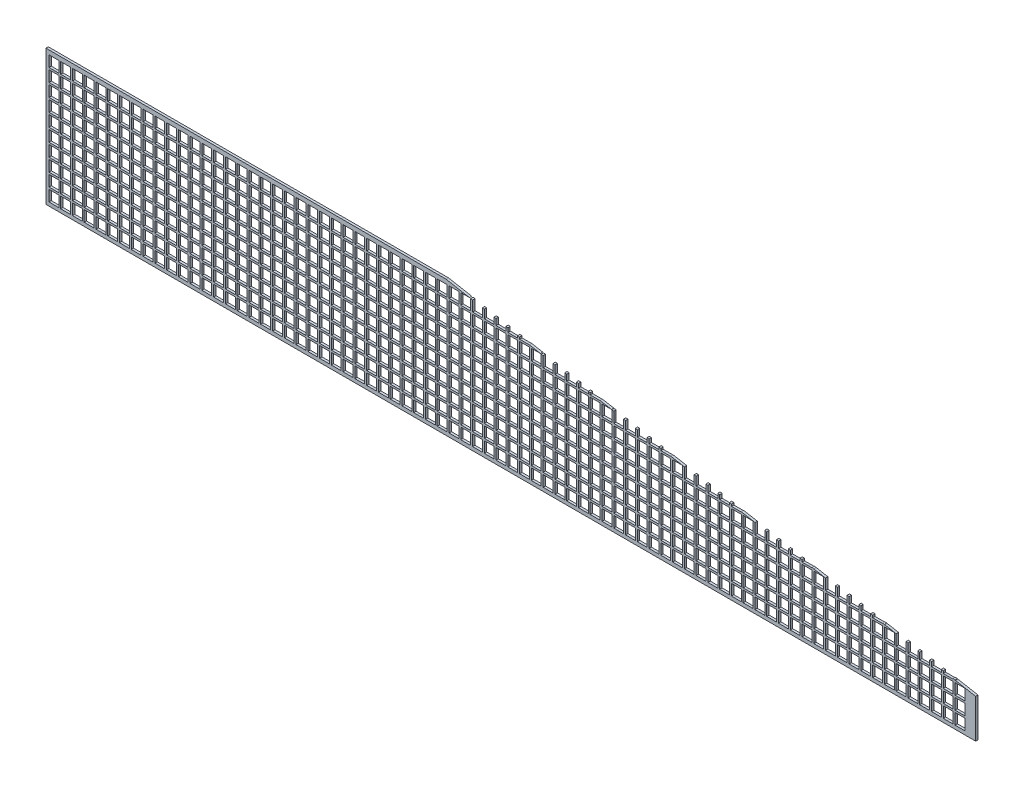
SolidWorks part; units mm, degrees
ref_plane "Front Plane" through (0, 0, 0) normal (0, 0, 1) x (1, 0, 0)
ref_plane "Top Plane" through (0, 0, 0) normal (0, 1, 0) x (1, 0, 0)
ref_plane "Right Plane" through (0, 0, 0) normal (1, 0, 0) x (0, 0, -1)
sketch "Sketch1" plane through (0, 0, 0) normal (0, 0, 1) x (1, 0, 0)
  line L1 (0, 0) -> (1003.3, 0)
  line L2 (0, 0) -> (0, 146.05)
  line L3 (0, 146.05) -> (431.8, 146.05)
  line L5 (1003.3, 0) -> (1003.3, 41.91)
  line L6 (1003.3, 41.91) -> (431.8, 146.05)
  line L7 (15.842, 141.4678) -> (26.4749, 141.4678)
  line L8 (3.142, 141.4678) -> (13.7749, 141.4678)
  line L9 (3.142, 141.4678) -> (3.142, 129.6081)
  line L10 (3.142, 129.6081) -> (13.7749, 129.6081)
  line L11 (13.7749, 141.4678) -> (13.7749, 129.6081)
  line L12 (15.842, 141.4678) -> (15.842, 129.6081)
  line L13 (15.842, 129.6081) -> (26.4749, 129.6081)
  line L14 (26.4749, 141.4678) -> (26.4749, 129.6081)
  line L15 (28.542, 141.4678) -> (39.1749, 141.4678)
  line L16 (28.542, 141.4678) -> (28.542, 129.6081)
  line L17 (28.542, 129.6081) -> (39.1749, 129.6081)
  line L18 (39.1749, 141.4678) -> (39.1749, 129.6081)
  line L19 (41.242, 141.4678) -> (51.8749, 141.4678)
  line L20 (41.242, 141.4678) -> (41.242, 129.6081)
  line L21 (41.242, 129.6081) -> (51.8749, 129.6081)
  line L22 (51.8749, 141.4678) -> (51.8749, 129.6081)
  line L23 (53.942, 141.4678) -> (64.5749, 141.4678)
  line L24 (53.942, 141.4678) -> (53.942, 129.6081)
  line L25 (53.942, 129.6081) -> (64.5749, 129.6081)
  line L26 (64.5749, 141.4678) -> (64.5749, 129.6081)
  line L27 (66.642, 141.4678) -> (77.2749, 141.4678)
  line L28 (66.642, 141.4678) -> (66.642, 129.6081)
  line L29 (66.642, 129.6081) -> (77.2749, 129.6081)
  line L30 (77.2749, 141.4678) -> (77.2749, 129.6081)
  line L31 (79.342, 141.4678) -> (89.9749, 141.4678)
  line L32 (79.342, 141.4678) -> (79.342, 129.6081)
  line L33 (79.342, 129.6081) -> (89.9749, 129.6081)
  line L34 (89.9749, 141.4678) -> (89.9749, 129.6081)
  line L35 (92.042, 141.4678) -> (102.6749, 141.4678)
  line L36 (92.042, 141.4678) -> (92.042, 129.6081)
  line L37 (92.042, 129.6081) -> (102.6749, 129.6081)
  line L38 (102.6749, 141.4678) -> (102.6749, 129.6081)
  line L39 (104.742, 141.4678) -> (115.3749, 141.4678)
  line L40 (104.742, 141.4678) -> (104.742, 129.6081)
  line L41 (104.742, 129.6081) -> (115.3749, 129.6081)
  line L42 (115.3749, 141.4678) -> (115.3749, 129.6081)
  line L43 (117.442, 141.4678) -> (128.0749, 141.4678)
  line L44 (117.442, 141.4678) -> (117.442, 129.6081)
  line L45 (117.442, 129.6081) -> (128.0749, 129.6081)
  line L46 (128.0749, 141.4678) -> (128.0749, 129.6081)
  line L47 (130.142, 141.4678) -> (140.7749, 141.4678)
  line L48 (130.142, 141.4678) -> (130.142, 129.6081)
  line L49 (130.142, 129.6081) -> (140.7749, 129.6081)
  line L50 (140.7749, 141.4678) -> (140.7749, 129.6081)
  line L51 (142.842, 141.4678) -> (153.4749, 141.4678)
  line L52 (142.842, 141.4678) -> (142.842, 129.6081)
  line L53 (142.842, 129.6081) -> (153.4749, 129.6081)
  line L54 (153.4749, 141.4678) -> (153.4749, 129.6081)
  line L55 (155.542, 141.4678) -> (166.1749, 141.4678)
  line L56 (155.542, 141.4678) -> (155.542, 129.6081)
  line L57 (155.542, 129.6081) -> (166.1749, 129.6081)
  line L58 (166.1749, 141.4678) -> (166.1749, 129.6081)
  line L59 (168.242, 141.4678) -> (178.8749, 141.4678)
  line L60 (168.242, 141.4678) -> (168.242, 129.6081)
  line L61 (168.242, 129.6081) -> (178.8749, 129.6081)
  line L62 (178.8749, 141.4678) -> (178.8749, 129.6081)
  line L63 (180.942, 141.4678) -> (191.5749, 141.4678)
  line L64 (180.942, 141.4678) -> (180.942, 129.6081)
  line L65 (180.942, 129.6081) -> (191.5749, 129.6081)
  line L66 (191.5749, 141.4678) -> (191.5749, 129.6081)
  line L67 (193.642, 141.4678) -> (204.2749, 141.4678)
  line L68 (193.642, 141.4678) -> (193.642, 129.6081)
  line L69 (193.642, 129.6081) -> (204.2749, 129.6081)
  line L70 (204.2749, 141.4678) -> (204.2749, 129.6081)
  line L71 (206.342, 141.4678) -> (216.9749, 141.4678)
  line L72 (206.342, 141.4678) -> (206.342, 129.6081)
  line L73 (206.342, 129.6081) -> (216.9749, 129.6081)
  line L74 (216.9749, 141.4678) -> (216.9749, 129.6081)
  line L75 (219.042, 141.4678) -> (229.6749, 141.4678)
  line L76 (219.042, 141.4678) -> (219.042, 129.6081)
  line L77 (219.042, 129.6081) -> (229.6749, 129.6081)
  line L78 (229.6749, 141.4678) -> (229.6749, 129.6081)
  line L79 (231.742, 141.4678) -> (242.3749, 141.4678)
  line L80 (231.742, 141.4678) -> (231.742, 129.6081)
  line L81 (231.742, 129.6081) -> (242.3749, 129.6081)
  line L82 (242.3749, 141.4678) -> (242.3749, 129.6081)
  line L83 (244.442, 141.4678) -> (255.0749, 141.4678)
  line L84 (244.442, 141.4678) -> (244.442, 129.6081)
  line L85 (244.442, 129.6081) -> (255.0749, 129.6081)
  line L86 (255.0749, 141.4678) -> (255.0749, 129.6081)
  line L87 (257.142, 141.4678) -> (267.7749, 141.4678)
  line L88 (257.142, 141.4678) -> (257.142, 129.6081)
  line L89 (257.142, 129.6081) -> (267.7749, 129.6081)
  line L90 (267.7749, 141.4678) -> (267.7749, 129.6081)
  line L91 (269.842, 141.4678) -> (280.4749, 141.4678)
  line L92 (269.842, 141.4678) -> (269.842, 129.6081)
  line L93 (269.842, 129.6081) -> (280.4749, 129.6081)
  line L94 (280.4749, 141.4678) -> (280.4749, 129.6081)
  line L95 (282.542, 141.4678) -> (293.1749, 141.4678)
  line L96 (282.542, 141.4678) -> (282.542, 129.6081)
  line L97 (282.542, 129.6081) -> (293.1749, 129.6081)
  line L98 (293.1749, 141.4678) -> (293.1749, 129.6081)
  line L99 (295.242, 141.4678) -> (305.8749, 141.4678)
  line L100 (295.242, 141.4678) -> (295.242, 129.6081)
  line L101 (295.242, 129.6081) -> (305.8749, 129.6081)
  line L102 (305.8749, 141.4678) -> (305.8749, 129.6081)
  line L103 (307.942, 141.4678) -> (318.5749, 141.4678)
  line L104 (307.942, 141.4678) -> (307.942, 129.6081)
  line L105 (307.942, 129.6081) -> (318.5749, 129.6081)
  line L106 (318.5749, 141.4678) -> (318.5749, 129.6081)
  line L107 (320.642, 141.4678) -> (331.2749, 141.4678)
  line L108 (320.642, 141.4678) -> (320.642, 129.6081)
  line L109 (320.642, 129.6081) -> (331.2749, 129.6081)
  line L110 (331.2749, 141.4678) -> (331.2749, 129.6081)
  line L111 (333.342, 141.4678) -> (343.9749, 141.4678)
  line L112 (333.342, 141.4678) -> (333.342, 129.6081)
  line L113 (333.342, 129.6081) -> (343.9749, 129.6081)
  line L114 (343.9749, 141.4678) -> (343.9749, 129.6081)
  line L115 (346.042, 141.4678) -> (356.6749, 141.4678)
  line L116 (346.042, 141.4678) -> (346.042, 129.6081)
  line L117 (346.042, 129.6081) -> (356.6749, 129.6081)
  line L118 (356.6749, 141.4678) -> (356.6749, 129.6081)
  line L119 (358.742, 141.4678) -> (369.3749, 141.4678)
  line L120 (358.742, 141.4678) -> (358.742, 129.6081)
  line L121 (358.742, 129.6081) -> (369.3749, 129.6081)
  line L122 (369.3749, 141.4678) -> (369.3749, 129.6081)
  line L123 (371.442, 141.4678) -> (382.0749, 141.4678)
  line L124 (371.442, 141.4678) -> (371.442, 129.6081)
  line L125 (371.442, 129.6081) -> (382.0749, 129.6081)
  line L126 (382.0749, 141.4678) -> (382.0749, 129.6081)
  line L127 (384.142, 141.4678) -> (394.7749, 141.4678)
  line L128 (384.142, 141.4678) -> (384.142, 129.6081)
  line L129 (384.142, 129.6081) -> (394.7749, 129.6081)
  line L130 (394.7749, 141.4678) -> (394.7749, 129.6081)
  line L131 (396.842, 141.4678) -> (407.4749, 141.4678)
  line L132 (396.842, 141.4678) -> (396.842, 129.6081)
  line L133 (396.842, 129.6081) -> (407.4749, 129.6081)
  line L134 (407.4749, 141.4678) -> (407.4749, 129.6081)
  line L135 (409.542, 141.4678) -> (420.1749, 141.4678)
  line L136 (409.542, 141.4678) -> (409.542, 129.6081)
  line L137 (409.542, 129.6081) -> (420.1749, 129.6081)
  line L138 (420.1749, 141.4678) -> (420.1749, 129.6081)
  line L139 (422.242, 141.4678) -> (432.8749, 141.4678)
  line L140 (422.242, 141.4678) -> (422.242, 129.6081)
  line L141 (422.242, 129.6081) -> (432.8749, 129.6081)
  line L142 (432.8749, 141.4678) -> (432.8749, 129.6081)
  line L143 (434.942, 141.4678) -> (445.5749, 141.4678)
  line L144 (434.942, 141.4678) -> (434.942, 129.6081)
  line L145 (434.942, 129.6081) -> (445.5749, 129.6081)
  line L146 (445.5749, 141.4678) -> (445.5749, 129.6081)
  line L147 (447.642, 141.4678) -> (458.2749, 141.4678)
  line L148 (447.642, 141.4678) -> (447.642, 129.6081)
  line L149 (447.642, 129.6081) -> (458.2749, 129.6081)
  line L150 (458.2749, 141.4678) -> (458.2749, 129.6081)
  line L151 (460.342, 141.4678) -> (470.9749, 141.4678)
  line L152 (460.342, 141.4678) -> (460.342, 129.6081)
  line L153 (460.342, 129.6081) -> (470.9749, 129.6081)
  line L154 (470.9749, 141.4678) -> (470.9749, 129.6081)
  line L155 (473.042, 141.4678) -> (483.6749, 141.4678)
  line L156 (473.042, 141.4678) -> (473.042, 129.6081)
  line L157 (473.042, 129.6081) -> (483.6749, 129.6081)
  line L158 (483.6749, 141.4678) -> (483.6749, 129.6081)
  line L159 (485.742, 141.4678) -> (496.3749, 141.4678)
  line L160 (485.742, 141.4678) -> (485.742, 129.6081)
  line L161 (485.742, 129.6081) -> (496.3749, 129.6081)
  line L162 (496.3749, 141.4678) -> (496.3749, 129.6081)
  line L163 (498.442, 141.4678) -> (509.0749, 141.4678)
  line L164 (498.442, 141.4678) -> (498.442, 129.6081)
  line L165 (498.442, 129.6081) -> (509.0749, 129.6081)
  line L166 (509.0749, 141.4678) -> (509.0749, 129.6081)
  line L167 (511.142, 141.4678) -> (521.7749, 141.4678)
  line L168 (511.142, 141.4678) -> (511.142, 129.6081)
  line L169 (511.142, 129.6081) -> (521.7749, 129.6081)
  line L170 (521.7749, 141.4678) -> (521.7749, 129.6081)
  line L171 (523.842, 141.4678) -> (534.4749, 141.4678)
  line L172 (523.842, 141.4678) -> (523.842, 129.6081)
  line L173 (523.842, 129.6081) -> (534.4749, 129.6081)
  line L174 (534.4749, 141.4678) -> (534.4749, 129.6081)
  line L175 (536.542, 141.4678) -> (547.1749, 141.4678)
  line L176 (536.542, 141.4678) -> (536.542, 129.6081)
  line L177 (536.542, 129.6081) -> (547.1749, 129.6081)
  line L178 (547.1749, 141.4678) -> (547.1749, 129.6081)
  line L179 (549.242, 141.4678) -> (559.8749, 141.4678)
  line L180 (549.242, 141.4678) -> (549.242, 129.6081)
  line L181 (549.242, 129.6081) -> (559.8749, 129.6081)
  line L182 (559.8749, 141.4678) -> (559.8749, 129.6081)
  line L183 (561.942, 141.4678) -> (572.5749, 141.4678)
  line L184 (561.942, 141.4678) -> (561.942, 129.6081)
  line L185 (561.942, 129.6081) -> (572.5749, 129.6081)
  line L186 (572.5749, 141.4678) -> (572.5749, 129.6081)
  line L187 (574.642, 141.4678) -> (585.2749, 141.4678)
  line L188 (574.642, 141.4678) -> (574.642, 129.6081)
  line L189 (574.642, 129.6081) -> (585.2749, 129.6081)
  line L190 (585.2749, 141.4678) -> (585.2749, 129.6081)
  line L191 (587.342, 141.4678) -> (597.9749, 141.4678)
  line L192 (587.342, 141.4678) -> (587.342, 129.6081)
  line L193 (587.342, 129.6081) -> (597.9749, 129.6081)
  line L194 (597.9749, 141.4678) -> (597.9749, 129.6081)
  line L195 (600.042, 141.4678) -> (610.6749, 141.4678)
  line L196 (600.042, 141.4678) -> (600.042, 129.6081)
  line L197 (600.042, 129.6081) -> (610.6749, 129.6081)
  line L198 (610.6749, 141.4678) -> (610.6749, 129.6081)
  line L199 (612.742, 141.4678) -> (623.3749, 141.4678)
  line L200 (612.742, 141.4678) -> (612.742, 129.6081)
  line L201 (612.742, 129.6081) -> (623.3749, 129.6081)
  line L202 (623.3749, 141.4678) -> (623.3749, 129.6081)
  line L203 (625.442, 141.4678) -> (636.0749, 141.4678)
  line L204 (625.442, 141.4678) -> (625.442, 129.6081)
  line L205 (625.442, 129.6081) -> (636.0749, 129.6081)
  line L206 (636.0749, 141.4678) -> (636.0749, 129.6081)
  line L207 (638.142, 141.4678) -> (648.7749, 141.4678)
  line L208 (638.142, 141.4678) -> (638.142, 129.6081)
  line L209 (638.142, 129.6081) -> (648.7749, 129.6081)
  line L210 (648.7749, 141.4678) -> (648.7749, 129.6081)
  line L211 (650.842, 141.4678) -> (661.4749, 141.4678)
  line L212 (650.842, 141.4678) -> (650.842, 129.6081)
  line L213 (650.842, 129.6081) -> (661.4749, 129.6081)
  line L214 (661.4749, 141.4678) -> (661.4749, 129.6081)
  line L215 (663.542, 141.4678) -> (674.1749, 141.4678)
  line L216 (663.542, 141.4678) -> (663.542, 129.6081)
  line L217 (663.542, 129.6081) -> (674.1749, 129.6081)
  line L218 (674.1749, 141.4678) -> (674.1749, 129.6081)
  line L219 (676.242, 141.4678) -> (686.8749, 141.4678)
  line L220 (676.242, 141.4678) -> (676.242, 129.6081)
  line L221 (676.242, 129.6081) -> (686.8749, 129.6081)
  line L222 (686.8749, 141.4678) -> (686.8749, 129.6081)
  line L223 (688.942, 141.4678) -> (699.5749, 141.4678)
  line L224 (688.942, 141.4678) -> (688.942, 129.6081)
  line L225 (688.942, 129.6081) -> (699.5749, 129.6081)
  line L226 (699.5749, 141.4678) -> (699.5749, 129.6081)
  line L227 (701.642, 141.4678) -> (712.2749, 141.4678)
  line L228 (701.642, 141.4678) -> (701.642, 129.6081)
  line L229 (701.642, 129.6081) -> (712.2749, 129.6081)
  line L230 (712.2749, 141.4678) -> (712.2749, 129.6081)
  line L231 (714.342, 141.4678) -> (724.9749, 141.4678)
  line L232 (714.342, 141.4678) -> (714.342, 129.6081)
  line L233 (714.342, 129.6081) -> (724.9749, 129.6081)
  line L234 (724.9749, 141.4678) -> (724.9749, 129.6081)
  line L235 (727.042, 141.4678) -> (737.6749, 141.4678)
  line L236 (727.042, 141.4678) -> (727.042, 129.6081)
  line L237 (727.042, 129.6081) -> (737.6749, 129.6081)
  line L238 (737.6749, 141.4678) -> (737.6749, 129.6081)
  line L239 (739.742, 141.4678) -> (750.3749, 141.4678)
  line L240 (739.742, 141.4678) -> (739.742, 129.6081)
  line L241 (739.742, 129.6081) -> (750.3749, 129.6081)
  line L242 (750.3749, 141.4678) -> (750.3749, 129.6081)
  line L243 (752.442, 141.4678) -> (763.0749, 141.4678)
  line L244 (752.442, 141.4678) -> (752.442, 129.6081)
  line L245 (752.442, 129.6081) -> (763.0749, 129.6081)
  line L246 (763.0749, 141.4678) -> (763.0749, 129.6081)
  line L247 (765.142, 141.4678) -> (775.7749, 141.4678)
  line L248 (765.142, 141.4678) -> (765.142, 129.6081)
  line L249 (765.142, 129.6081) -> (775.7749, 129.6081)
  line L250 (775.7749, 141.4678) -> (775.7749, 129.6081)
  line L251 (777.842, 141.4678) -> (788.4749, 141.4678)
  line L252 (777.842, 141.4678) -> (777.842, 129.6081)
  line L253 (777.842, 129.6081) -> (788.4749, 129.6081)
  line L254 (788.4749, 141.4678) -> (788.4749, 129.6081)
  line L255 (790.542, 141.4678) -> (801.1749, 141.4678)
  line L256 (790.542, 141.4678) -> (790.542, 129.6081)
  line L257 (790.542, 129.6081) -> (801.1749, 129.6081)
  line L258 (801.1749, 141.4678) -> (801.1749, 129.6081)
  line L259 (803.242, 141.4678) -> (813.8749, 141.4678)
  line L260 (803.242, 141.4678) -> (803.242, 129.6081)
  line L261 (803.242, 129.6081) -> (813.8749, 129.6081)
  line L262 (813.8749, 141.4678) -> (813.8749, 129.6081)
  line L263 (815.942, 141.4678) -> (826.5749, 141.4678)
  line L264 (815.942, 141.4678) -> (815.942, 129.6081)
  line L265 (815.942, 129.6081) -> (826.5749, 129.6081)
  line L266 (826.5749, 141.4678) -> (826.5749, 129.6081)
  line L267 (828.642, 141.4678) -> (839.2749, 141.4678)
  line L268 (828.642, 141.4678) -> (828.642, 129.6081)
  line L269 (828.642, 129.6081) -> (839.2749, 129.6081)
  line L270 (839.2749, 141.4678) -> (839.2749, 129.6081)
  line L271 (841.342, 141.4678) -> (851.9749, 141.4678)
  line L272 (841.342, 141.4678) -> (841.342, 129.6081)
  line L273 (841.342, 129.6081) -> (851.9749, 129.6081)
  line L274 (851.9749, 141.4678) -> (851.9749, 129.6081)
  line L275 (854.042, 141.4678) -> (864.6749, 141.4678)
  line L276 (854.042, 141.4678) -> (854.042, 129.6081)
  line L277 (854.042, 129.6081) -> (864.6749, 129.6081)
  line L278 (864.6749, 141.4678) -> (864.6749, 129.6081)
  line L279 (866.742, 141.4678) -> (877.3749, 141.4678)
  line L280 (866.742, 141.4678) -> (866.742, 129.6081)
  line L281 (866.742, 129.6081) -> (877.3749, 129.6081)
  line L282 (877.3749, 141.4678) -> (877.3749, 129.6081)
  line L283 (879.442, 141.4678) -> (890.0749, 141.4678)
  line L284 (879.442, 141.4678) -> (879.442, 129.6081)
  line L285 (879.442, 129.6081) -> (890.0749, 129.6081)
  line L286 (890.0749, 141.4678) -> (890.0749, 129.6081)
  line L287 (892.142, 141.4678) -> (902.7749, 141.4678)
  line L288 (892.142, 141.4678) -> (892.142, 129.6081)
  line L289 (892.142, 129.6081) -> (902.7749, 129.6081)
  line L290 (902.7749, 141.4678) -> (902.7749, 129.6081)
  line L291 (904.842, 141.4678) -> (915.4749, 141.4678)
  line L292 (904.842, 141.4678) -> (904.842, 129.6081)
  line L293 (904.842, 129.6081) -> (915.4749, 129.6081)
  line L294 (915.4749, 141.4678) -> (915.4749, 129.6081)
  line L295 (917.542, 141.4678) -> (928.1749, 141.4678)
  line L296 (917.542, 141.4678) -> (917.542, 129.6081)
  line L297 (917.542, 129.6081) -> (928.1749, 129.6081)
  line L298 (928.1749, 141.4678) -> (928.1749, 129.6081)
  line L299 (930.242, 141.4678) -> (940.8749, 141.4678)
  line L300 (930.242, 141.4678) -> (930.242, 129.6081)
  line L301 (930.242, 129.6081) -> (940.8749, 129.6081)
  line L302 (940.8749, 141.4678) -> (940.8749, 129.6081)
  line L303 (942.942, 141.4678) -> (953.5749, 141.4678)
  line L304 (942.942, 141.4678) -> (942.942, 129.6081)
  line L305 (942.942, 129.6081) -> (953.5749, 129.6081)
  line L306 (953.5749, 141.4678) -> (953.5749, 129.6081)
  line L307 (955.642, 141.4678) -> (966.2749, 141.4678)
  line L308 (955.642, 141.4678) -> (955.642, 129.6081)
  line L309 (955.642, 129.6081) -> (966.2749, 129.6081)
  line L310 (966.2749, 141.4678) -> (966.2749, 129.6081)
  line L311 (968.342, 141.4678) -> (978.9749, 141.4678)
  line L312 (968.342, 141.4678) -> (968.342, 129.6081)
  line L313 (968.342, 129.6081) -> (978.9749, 129.6081)
  line L314 (978.9749, 141.4678) -> (978.9749, 129.6081)
  line L315 (981.042, 141.4678) -> (991.6749, 141.4678)
  line L316 (981.042, 141.4678) -> (981.042, 129.6081)
  line L317 (981.042, 129.6081) -> (991.6749, 129.6081)
  line L318 (991.6749, 141.4678) -> (991.6749, 129.6081)
  line L319 (15.842, 127.4978) -> (26.4749, 127.4978)
  line L320 (15.842, 127.4978) -> (15.842, 115.6381)
  line L321 (15.842, 115.6381) -> (26.4749, 115.6381)
  line L322 (26.4749, 127.4978) -> (26.4749, 115.6381)
  line L323 (28.542, 127.4978) -> (39.1749, 127.4978)
  line L324 (28.542, 127.4978) -> (28.542, 115.6381)
  line L325 (28.542, 115.6381) -> (39.1749, 115.6381)
  line L326 (39.1749, 127.4978) -> (39.1749, 115.6381)
  line L327 (41.242, 127.4978) -> (51.8749, 127.4978)
  line L328 (41.242, 127.4978) -> (41.242, 115.6381)
  line L329 (41.242, 115.6381) -> (51.8749, 115.6381)
  line L330 (51.8749, 127.4978) -> (51.8749, 115.6381)
  line L331 (53.942, 127.4978) -> (64.5749, 127.4978)
  line L332 (53.942, 127.4978) -> (53.942, 115.6381)
  line L333 (53.942, 115.6381) -> (64.5749, 115.6381)
  line L334 (64.5749, 127.4978) -> (64.5749, 115.6381)
  line L335 (66.642, 127.4978) -> (77.2749, 127.4978)
  line L336 (66.642, 127.4978) -> (66.642, 115.6381)
  line L337 (66.642, 115.6381) -> (77.2749, 115.6381)
  line L338 (77.2749, 127.4978) -> (77.2749, 115.6381)
  line L339 (79.342, 127.4978) -> (89.9749, 127.4978)
  line L340 (79.342, 127.4978) -> (79.342, 115.6381)
  line L341 (79.342, 115.6381) -> (89.9749, 115.6381)
  line L342 (89.9749, 127.4978) -> (89.9749, 115.6381)
  line L343 (92.042, 127.4978) -> (102.6749, 127.4978)
  line L344 (92.042, 127.4978) -> (92.042, 115.6381)
  line L345 (92.042, 115.6381) -> (102.6749, 115.6381)
  line L346 (102.6749, 127.4978) -> (102.6749, 115.6381)
  line L347 (104.742, 127.4978) -> (115.3749, 127.4978)
  line L348 (104.742, 127.4978) -> (104.742, 115.6381)
  line L349 (104.742, 115.6381) -> (115.3749, 115.6381)
  line L350 (115.3749, 127.4978) -> (115.3749, 115.6381)
  line L351 (117.442, 127.4978) -> (128.0749, 127.4978)
  line L352 (117.442, 127.4978) -> (117.442, 115.6381)
  line L353 (117.442, 115.6381) -> (128.0749, 115.6381)
  line L354 (128.0749, 127.4978) -> (128.0749, 115.6381)
  line L355 (130.142, 127.4978) -> (140.7749, 127.4978)
  line L356 (130.142, 127.4978) -> (130.142, 115.6381)
  line L357 (130.142, 115.6381) -> (140.7749, 115.6381)
  line L358 (140.7749, 127.4978) -> (140.7749, 115.6381)
  line L359 (142.842, 127.4978) -> (153.4749, 127.4978)
  line L360 (142.842, 127.4978) -> (142.842, 115.6381)
  line L361 (142.842, 115.6381) -> (153.4749, 115.6381)
  line L362 (153.4749, 127.4978) -> (153.4749, 115.6381)
  line L363 (155.542, 127.4978) -> (166.1749, 127.4978)
  line L364 (155.542, 127.4978) -> (155.542, 115.6381)
  line L365 (155.542, 115.6381) -> (166.1749, 115.6381)
  line L366 (166.1749, 127.4978) -> (166.1749, 115.6381)
  line L367 (168.242, 127.4978) -> (178.8749, 127.4978)
  line L368 (168.242, 127.4978) -> (168.242, 115.6381)
  line L369 (168.242, 115.6381) -> (178.8749, 115.6381)
  line L370 (178.8749, 127.4978) -> (178.8749, 115.6381)
  line L371 (180.942, 127.4978) -> (191.5749, 127.4978)
  line L372 (180.942, 127.4978) -> (180.942, 115.6381)
  line L373 (180.942, 115.6381) -> (191.5749, 115.6381)
  line L374 (191.5749, 127.4978) -> (191.5749, 115.6381)
  line L375 (193.642, 127.4978) -> (204.2749, 127.4978)
  line L376 (193.642, 127.4978) -> (193.642, 115.6381)
  line L377 (193.642, 115.6381) -> (204.2749, 115.6381)
  line L378 (204.2749, 127.4978) -> (204.2749, 115.6381)
  line L379 (206.342, 127.4978) -> (216.9749, 127.4978)
  line L380 (206.342, 127.4978) -> (206.342, 115.6381)
  line L381 (206.342, 115.6381) -> (216.9749, 115.6381)
  line L382 (216.9749, 127.4978) -> (216.9749, 115.6381)
  line L383 (219.042, 127.4978) -> (229.6749, 127.4978)
  line L384 (219.042, 127.4978) -> (219.042, 115.6381)
  line L385 (219.042, 115.6381) -> (229.6749, 115.6381)
  line L386 (229.6749, 127.4978) -> (229.6749, 115.6381)
  line L387 (231.742, 127.4978) -> (242.3749, 127.4978)
  line L388 (231.742, 127.4978) -> (231.742, 115.6381)
  line L389 (231.742, 115.6381) -> (242.3749, 115.6381)
  line L390 (242.3749, 127.4978) -> (242.3749, 115.6381)
  line L391 (244.442, 127.4978) -> (255.0749, 127.4978)
  line L392 (244.442, 127.4978) -> (244.442, 115.6381)
  line L393 (244.442, 115.6381) -> (255.0749, 115.6381)
  line L394 (255.0749, 127.4978) -> (255.0749, 115.6381)
  line L395 (257.142, 127.4978) -> (267.7749, 127.4978)
  line L396 (257.142, 127.4978) -> (257.142, 115.6381)
  line L397 (257.142, 115.6381) -> (267.7749, 115.6381)
  line L398 (267.7749, 127.4978) -> (267.7749, 115.6381)
  line L399 (269.842, 127.4978) -> (280.4749, 127.4978)
  line L400 (269.842, 127.4978) -> (269.842, 115.6381)
  line L401 (269.842, 115.6381) -> (280.4749, 115.6381)
  line L402 (280.4749, 127.4978) -> (280.4749, 115.6381)
  line L403 (282.542, 127.4978) -> (293.1749, 127.4978)
  line L404 (282.542, 127.4978) -> (282.542, 115.6381)
  line L405 (282.542, 115.6381) -> (293.1749, 115.6381)
  line L406 (293.1749, 127.4978) -> (293.1749, 115.6381)
  line L407 (295.242, 127.4978) -> (305.8749, 127.4978)
  line L408 (295.242, 127.4978) -> (295.242, 115.6381)
  line L409 (295.242, 115.6381) -> (305.8749, 115.6381)
  line L410 (305.8749, 127.4978) -> (305.8749, 115.6381)
  line L411 (307.942, 127.4978) -> (318.5749, 127.4978)
  line L412 (307.942, 127.4978) -> (307.942, 115.6381)
  line L413 (307.942, 115.6381) -> (318.5749, 115.6381)
  line L414 (318.5749, 127.4978) -> (318.5749, 115.6381)
  line L415 (320.642, 127.4978) -> (331.2749, 127.4978)
  line L416 (320.642, 127.4978) -> (320.642, 115.6381)
  line L417 (320.642, 115.6381) -> (331.2749, 115.6381)
  line L418 (331.2749, 127.4978) -> (331.2749, 115.6381)
  line L419 (333.342, 127.4978) -> (343.9749, 127.4978)
  line L420 (333.342, 127.4978) -> (333.342, 115.6381)
  line L421 (333.342, 115.6381) -> (343.9749, 115.6381)
  line L422 (343.9749, 127.4978) -> (343.9749, 115.6381)
  line L423 (346.042, 127.4978) -> (356.6749, 127.4978)
  line L424 (346.042, 127.4978) -> (346.042, 115.6381)
  line L425 (346.042, 115.6381) -> (356.6749, 115.6381)
  line L426 (356.6749, 127.4978) -> (356.6749, 115.6381)
  line L427 (358.742, 127.4978) -> (369.3749, 127.4978)
  line L428 (358.742, 127.4978) -> (358.742, 115.6381)
  line L429 (358.742, 115.6381) -> (369.3749, 115.6381)
  line L430 (369.3749, 127.4978) -> (369.3749, 115.6381)
  line L431 (371.442, 127.4978) -> (382.0749, 127.4978)
  line L432 (371.442, 127.4978) -> (371.442, 115.6381)
  line L433 (371.442, 115.6381) -> (382.0749, 115.6381)
  line L434 (382.0749, 127.4978) -> (382.0749, 115.6381)
  line L435 (384.142, 127.4978) -> (394.7749, 127.4978)
  line L436 (384.142, 127.4978) -> (384.142, 115.6381)
  line L437 (384.142, 115.6381) -> (394.7749, 115.6381)
  line L438 (394.7749, 127.4978) -> (394.7749, 115.6381)
  line L439 (396.842, 127.4978) -> (407.4749, 127.4978)
  line L440 (396.842, 127.4978) -> (396.842, 115.6381)
  line L441 (396.842, 115.6381) -> (407.4749, 115.6381)
  line L442 (407.4749, 127.4978) -> (407.4749, 115.6381)
  line L443 (409.542, 127.4978) -> (420.1749, 127.4978)
  line L444 (409.542, 127.4978) -> (409.542, 115.6381)
  line L445 (409.542, 115.6381) -> (420.1749, 115.6381)
  line L446 (420.1749, 127.4978) -> (420.1749, 115.6381)
  line L447 (422.242, 127.4978) -> (432.8749, 127.4978)
  line L448 (422.242, 127.4978) -> (422.242, 115.6381)
  line L449 (422.242, 115.6381) -> (432.8749, 115.6381)
  line L450 (432.8749, 127.4978) -> (432.8749, 115.6381)
  line L451 (434.942, 127.4978) -> (445.5749, 127.4978)
  line L452 (434.942, 127.4978) -> (434.942, 115.6381)
  line L453 (434.942, 115.6381) -> (445.5749, 115.6381)
  line L454 (445.5749, 127.4978) -> (445.5749, 115.6381)
  line L455 (447.642, 127.4978) -> (458.2749, 127.4978)
  line L456 (447.642, 127.4978) -> (447.642, 115.6381)
  line L457 (447.642, 115.6381) -> (458.2749, 115.6381)
  line L458 (458.2749, 127.4978) -> (458.2749, 115.6381)
  line L459 (460.342, 127.4978) -> (470.9749, 127.4978)
  line L460 (460.342, 127.4978) -> (460.342, 115.6381)
  line L461 (460.342, 115.6381) -> (470.9749, 115.6381)
  line L462 (470.9749, 127.4978) -> (470.9749, 115.6381)
  line L463 (473.042, 127.4978) -> (483.6749, 127.4978)
  line L464 (473.042, 127.4978) -> (473.042, 115.6381)
  line L465 (473.042, 115.6381) -> (483.6749, 115.6381)
  line L466 (483.6749, 127.4978) -> (483.6749, 115.6381)
  line L467 (485.742, 127.4978) -> (496.3749, 127.4978)
  line L468 (485.742, 127.4978) -> (485.742, 115.6381)
  line L469 (485.742, 115.6381) -> (496.3749, 115.6381)
  line L470 (496.3749, 127.4978) -> (496.3749, 115.6381)
  line L471 (498.442, 127.4978) -> (509.0749, 127.4978)
  line L472 (498.442, 127.4978) -> (498.442, 115.6381)
  line L473 (498.442, 115.6381) -> (509.0749, 115.6381)
  line L474 (509.0749, 127.4978) -> (509.0749, 115.6381)
  line L475 (511.142, 127.4978) -> (521.7749, 127.4978)
  line L476 (511.142, 127.4978) -> (511.142, 115.6381)
  line L477 (511.142, 115.6381) -> (521.7749, 115.6381)
  line L478 (521.7749, 127.4978) -> (521.7749, 115.6381)
  line L479 (523.842, 127.4978) -> (534.4749, 127.4978)
  line L480 (523.842, 127.4978) -> (523.842, 115.6381)
  line L481 (523.842, 115.6381) -> (534.4749, 115.6381)
  line L482 (534.4749, 127.4978) -> (534.4749, 115.6381)
  line L483 (536.542, 127.4978) -> (547.1749, 127.4978)
  line L484 (536.542, 127.4978) -> (536.542, 115.6381)
  line L485 (536.542, 115.6381) -> (547.1749, 115.6381)
  line L486 (547.1749, 127.4978) -> (547.1749, 115.6381)
  line L487 (549.242, 127.4978) -> (559.8749, 127.4978)
  line L488 (549.242, 127.4978) -> (549.242, 115.6381)
  line L489 (549.242, 115.6381) -> (559.8749, 115.6381)
  line L490 (559.8749, 127.4978) -> (559.8749, 115.6381)
  line L491 (561.942, 127.4978) -> (572.5749, 127.4978)
  line L492 (561.942, 127.4978) -> (561.942, 115.6381)
  line L493 (561.942, 115.6381) -> (572.5749, 115.6381)
  line L494 (572.5749, 127.4978) -> (572.5749, 115.6381)
  line L495 (574.642, 127.4978) -> (585.2749, 127.4978)
  line L496 (574.642, 127.4978) -> (574.642, 115.6381)
  line L497 (574.642, 115.6381) -> (585.2749, 115.6381)
  line L498 (585.2749, 127.4978) -> (585.2749, 115.6381)
  line L499 (587.342, 127.4978) -> (597.9749, 127.4978)
  line L500 (587.342, 127.4978) -> (587.342, 115.6381)
  line L501 (587.342, 115.6381) -> (597.9749, 115.6381)
  line L502 (597.9749, 127.4978) -> (597.9749, 115.6381)
  line L503 (600.042, 127.4978) -> (610.6749, 127.4978)
  line L504 (600.042, 127.4978) -> (600.042, 115.6381)
  line L505 (600.042, 115.6381) -> (610.6749, 115.6381)
  line L506 (610.6749, 127.4978) -> (610.6749, 115.6381)
  line L507 (612.742, 127.4978) -> (623.3749, 127.4978)
  line L508 (612.742, 127.4978) -> (612.742, 115.6381)
  line L509 (612.742, 115.6381) -> (623.3749, 115.6381)
  line L510 (623.3749, 127.4978) -> (623.3749, 115.6381)
  line L511 (625.442, 127.4978) -> (636.0749, 127.4978)
  line L512 (625.442, 127.4978) -> (625.442, 115.6381)
  line L513 (625.442, 115.6381) -> (636.0749, 115.6381)
  line L514 (636.0749, 127.4978) -> (636.0749, 115.6381)
  line L515 (638.142, 127.4978) -> (648.7749, 127.4978)
  line L516 (638.142, 127.4978) -> (638.142, 115.6381)
  line L517 (638.142, 115.6381) -> (648.7749, 115.6381)
  line L518 (648.7749, 127.4978) -> (648.7749, 115.6381)
  line L519 (650.842, 127.4978) -> (661.4749, 127.4978)
  line L520 (650.842, 127.4978) -> (650.842, 115.6381)
  line L521 (650.842, 115.6381) -> (661.4749, 115.6381)
  line L522 (661.4749, 127.4978) -> (661.4749, 115.6381)
  line L523 (663.542, 127.4978) -> (674.1749, 127.4978)
  line L524 (663.542, 127.4978) -> (663.542, 115.6381)
  line L525 (663.542, 115.6381) -> (674.1749, 115.6381)
  line L526 (674.1749, 127.4978) -> (674.1749, 115.6381)
  line L527 (676.242, 127.4978) -> (686.8749, 127.4978)
  line L528 (676.242, 127.4978) -> (676.242, 115.6381)
  line L529 (676.242, 115.6381) -> (686.8749, 115.6381)
  line L530 (686.8749, 127.4978) -> (686.8749, 115.6381)
  line L531 (688.942, 127.4978) -> (699.5749, 127.4978)
  line L532 (688.942, 127.4978) -> (688.942, 115.6381)
  line L533 (688.942, 115.6381) -> (699.5749, 115.6381)
  line L534 (699.5749, 127.4978) -> (699.5749, 115.6381)
  line L535 (701.642, 127.4978) -> (712.2749, 127.4978)
  line L536 (701.642, 127.4978) -> (701.642, 115.6381)
  line L537 (701.642, 115.6381) -> (712.2749, 115.6381)
  line L538 (712.2749, 127.4978) -> (712.2749, 115.6381)
  line L539 (714.342, 127.4978) -> (724.9749, 127.4978)
  line L540 (714.342, 127.4978) -> (714.342, 115.6381)
  line L541 (714.342, 115.6381) -> (724.9749, 115.6381)
  line L542 (724.9749, 127.4978) -> (724.9749, 115.6381)
  line L543 (727.042, 127.4978) -> (737.6749, 127.4978)
  line L544 (727.042, 127.4978) -> (727.042, 115.6381)
  line L545 (727.042, 115.6381) -> (737.6749, 115.6381)
  line L546 (737.6749, 127.4978) -> (737.6749, 115.6381)
  line L547 (739.742, 127.4978) -> (750.3749, 127.4978)
  line L548 (739.742, 127.4978) -> (739.742, 115.6381)
  line L549 (739.742, 115.6381) -> (750.3749, 115.6381)
  line L550 (750.3749, 127.4978) -> (750.3749, 115.6381)
  line L551 (752.442, 127.4978) -> (763.0749, 127.4978)
  line L552 (752.442, 127.4978) -> (752.442, 115.6381)
  line L553 (752.442, 115.6381) -> (763.0749, 115.6381)
  line L554 (763.0749, 127.4978) -> (763.0749, 115.6381)
  line L555 (765.142, 127.4978) -> (775.7749, 127.4978)
  line L556 (765.142, 127.4978) -> (765.142, 115.6381)
  line L557 (765.142, 115.6381) -> (775.7749, 115.6381)
  line L558 (775.7749, 127.4978) -> (775.7749, 115.6381)
  line L559 (777.842, 127.4978) -> (788.4749, 127.4978)
  line L560 (777.842, 127.4978) -> (777.842, 115.6381)
  line L561 (777.842, 115.6381) -> (788.4749, 115.6381)
  line L562 (788.4749, 127.4978) -> (788.4749, 115.6381)
  line L563 (790.542, 127.4978) -> (801.1749, 127.4978)
  line L564 (790.542, 127.4978) -> (790.542, 115.6381)
  line L565 (790.542, 115.6381) -> (801.1749, 115.6381)
  line L566 (801.1749, 127.4978) -> (801.1749, 115.6381)
  line L567 (803.242, 127.4978) -> (813.8749, 127.4978)
  line L568 (803.242, 127.4978) -> (803.242, 115.6381)
  line L569 (803.242, 115.6381) -> (813.8749, 115.6381)
  line L570 (813.8749, 127.4978) -> (813.8749, 115.6381)
  line L571 (815.942, 127.4978) -> (826.5749, 127.4978)
  line L572 (815.942, 127.4978) -> (815.942, 115.6381)
  line L573 (815.942, 115.6381) -> (826.5749, 115.6381)
  line L574 (826.5749, 127.4978) -> (826.5749, 115.6381)
  line L575 (828.642, 127.4978) -> (839.2749, 127.4978)
  line L576 (828.642, 127.4978) -> (828.642, 115.6381)
  line L577 (828.642, 115.6381) -> (839.2749, 115.6381)
  line L578 (839.2749, 127.4978) -> (839.2749, 115.6381)
  line L579 (841.342, 127.4978) -> (851.9749, 127.4978)
  line L580 (841.342, 127.4978) -> (841.342, 115.6381)
  line L581 (841.342, 115.6381) -> (851.9749, 115.6381)
  line L582 (851.9749, 127.4978) -> (851.9749, 115.6381)
  line L583 (854.042, 127.4978) -> (864.6749, 127.4978)
  line L584 (854.042, 127.4978) -> (854.042, 115.6381)
  line L585 (854.042, 115.6381) -> (864.6749, 115.6381)
  line L586 (864.6749, 127.4978) -> (864.6749, 115.6381)
  line L587 (866.742, 127.4978) -> (877.3749, 127.4978)
  line L588 (866.742, 127.4978) -> (866.742, 115.6381)
  line L589 (866.742, 115.6381) -> (877.3749, 115.6381)
  line L590 (877.3749, 127.4978) -> (877.3749, 115.6381)
  line L591 (879.442, 127.4978) -> (890.0749, 127.4978)
  line L592 (879.442, 127.4978) -> (879.442, 115.6381)
  line L593 (879.442, 115.6381) -> (890.0749, 115.6381)
  line L594 (890.0749, 127.4978) -> (890.0749, 115.6381)
  line L595 (892.142, 127.4978) -> (902.7749, 127.4978)
  line L596 (892.142, 127.4978) -> (892.142, 115.6381)
  line L597 (892.142, 115.6381) -> (902.7749, 115.6381)
  line L598 (902.7749, 127.4978) -> (902.7749, 115.6381)
  line L599 (904.842, 127.4978) -> (915.4749, 127.4978)
  line L600 (904.842, 127.4978) -> (904.842, 115.6381)
  line L601 (904.842, 115.6381) -> (915.4749, 115.6381)
  line L602 (915.4749, 127.4978) -> (915.4749, 115.6381)
  line L603 (917.542, 127.4978) -> (928.1749, 127.4978)
  line L604 (917.542, 127.4978) -> (917.542, 115.6381)
  line L605 (917.542, 115.6381) -> (928.1749, 115.6381)
  line L606 (928.1749, 127.4978) -> (928.1749, 115.6381)
  line L607 (930.242, 127.4978) -> (940.8749, 127.4978)
  line L608 (930.242, 127.4978) -> (930.242, 115.6381)
  line L609 (930.242, 115.6381) -> (940.8749, 115.6381)
  line L610 (940.8749, 127.4978) -> (940.8749, 115.6381)
  line L611 (942.942, 127.4978) -> (953.5749, 127.4978)
  line L612 (942.942, 127.4978) -> (942.942, 115.6381)
  line L613 (942.942, 115.6381) -> (953.5749, 115.6381)
  line L614 (953.5749, 127.4978) -> (953.5749, 115.6381)
  line L615 (955.642, 127.4978) -> (966.2749, 127.4978)
  line L616 (955.642, 127.4978) -> (955.642, 115.6381)
  line L617 (955.642, 115.6381) -> (966.2749, 115.6381)
  line L618 (966.2749, 127.4978) -> (966.2749, 115.6381)
  line L619 (968.342, 127.4978) -> (978.9749, 127.4978)
  line L620 (968.342, 127.4978) -> (968.342, 115.6381)
  line L621 (968.342, 115.6381) -> (978.9749, 115.6381)
  line L622 (978.9749, 127.4978) -> (978.9749, 115.6381)
  line L623 (981.042, 127.4978) -> (991.6749, 127.4978)
  line L624 (981.042, 127.4978) -> (981.042, 115.6381)
  line L625 (981.042, 115.6381) -> (991.6749, 115.6381)
  line L626 (991.6749, 127.4978) -> (991.6749, 115.6381)
  line L627 (15.842, 113.5278) -> (26.4749, 113.5278)
  line L628 (15.842, 113.5278) -> (15.842, 101.6681)
  line L629 (15.842, 101.6681) -> (26.4749, 101.6681)
  line L630 (26.4749, 113.5278) -> (26.4749, 101.6681)
  line L631 (28.542, 113.5278) -> (39.1749, 113.5278)
  line L632 (28.542, 113.5278) -> (28.542, 101.6681)
  line L633 (28.542, 101.6681) -> (39.1749, 101.6681)
  line L634 (39.1749, 113.5278) -> (39.1749, 101.6681)
  line L635 (41.242, 113.5278) -> (51.8749, 113.5278)
  line L636 (41.242, 113.5278) -> (41.242, 101.6681)
  line L637 (41.242, 101.6681) -> (51.8749, 101.6681)
  line L638 (51.8749, 113.5278) -> (51.8749, 101.6681)
  line L639 (53.942, 113.5278) -> (64.5749, 113.5278)
  line L640 (53.942, 113.5278) -> (53.942, 101.6681)
  line L641 (53.942, 101.6681) -> (64.5749, 101.6681)
  line L642 (64.5749, 113.5278) -> (64.5749, 101.6681)
  line L643 (66.642, 113.5278) -> (77.2749, 113.5278)
  line L644 (66.642, 113.5278) -> (66.642, 101.6681)
  line L645 (66.642, 101.6681) -> (77.2749, 101.6681)
  line L646 (77.2749, 113.5278) -> (77.2749, 101.6681)
  line L647 (79.342, 113.5278) -> (89.9749, 113.5278)
  line L648 (79.342, 113.5278) -> (79.342, 101.6681)
  line L649 (79.342, 101.6681) -> (89.9749, 101.6681)
  line L650 (89.9749, 113.5278) -> (89.9749, 101.6681)
  line L651 (92.042, 113.5278) -> (102.6749, 113.5278)
  line L652 (92.042, 113.5278) -> (92.042, 101.6681)
  line L653 (92.042, 101.6681) -> (102.6749, 101.6681)
  line L654 (102.6749, 113.5278) -> (102.6749, 101.6681)
  line L655 (104.742, 113.5278) -> (115.3749, 113.5278)
  line L656 (104.742, 113.5278) -> (104.742, 101.6681)
  line L657 (104.742, 101.6681) -> (115.3749, 101.6681)
  line L658 (115.3749, 113.5278) -> (115.3749, 101.6681)
  line L659 (117.442, 113.5278) -> (128.0749, 113.5278)
  line L660 (117.442, 113.5278) -> (117.442, 101.6681)
  line L661 (117.442, 101.6681) -> (128.0749, 101.6681)
  line L662 (128.0749, 113.5278) -> (128.0749, 101.6681)
  line L663 (130.142, 113.5278) -> (140.7749, 113.5278)
  line L664 (130.142, 113.5278) -> (130.142, 101.6681)
  line L665 (130.142, 101.6681) -> (140.7749, 101.6681)
  line L666 (140.7749, 113.5278) -> (140.7749, 101.6681)
  line L667 (142.842, 113.5278) -> (153.4749, 113.5278)
  line L668 (142.842, 113.5278) -> (142.842, 101.6681)
  line L669 (142.842, 101.6681) -> (153.4749, 101.6681)
  line L670 (153.4749, 113.5278) -> (153.4749, 101.6681)
  line L671 (155.542, 113.5278) -> (166.1749, 113.5278)
  line L672 (155.542, 113.5278) -> (155.542, 101.6681)
  line L673 (155.542, 101.6681) -> (166.1749, 101.6681)
  line L674 (166.1749, 113.5278) -> (166.1749, 101.6681)
  line L675 (168.242, 113.5278) -> (178.8749, 113.5278)
  line L676 (168.242, 113.5278) -> (168.242, 101.6681)
  line L677 (168.242, 101.6681) -> (178.8749, 101.6681)
  line L678 (178.8749, 113.5278) -> (178.8749, 101.6681)
  line L679 (180.942, 113.5278) -> (191.5749, 113.5278)
  line L680 (180.942, 113.5278) -> (180.942, 101.6681)
  line L681 (180.942, 101.6681) -> (191.5749, 101.6681)
  line L682 (191.5749, 113.5278) -> (191.5749, 101.6681)
  line L683 (193.642, 113.5278) -> (204.2749, 113.5278)
  line L684 (193.642, 113.5278) -> (193.642, 101.6681)
  line L685 (193.642, 101.6681) -> (204.2749, 101.6681)
  line L686 (204.2749, 113.5278) -> (204.2749, 101.6681)
  line L687 (206.342, 113.5278) -> (216.9749, 113.5278)
  line L688 (206.342, 113.5278) -> (206.342, 101.6681)
  line L689 (206.342, 101.6681) -> (216.9749, 101.6681)
  line L690 (216.9749, 113.5278) -> (216.9749, 101.6681)
  line L691 (219.042, 113.5278) -> (229.6749, 113.5278)
  line L692 (219.042, 113.5278) -> (219.042, 101.6681)
  line L693 (219.042, 101.6681) -> (229.6749, 101.6681)
  line L694 (229.6749, 113.5278) -> (229.6749, 101.6681)
  line L695 (231.742, 113.5278) -> (242.3749, 113.5278)
  line L696 (231.742, 113.5278) -> (231.742, 101.6681)
  line L697 (231.742, 101.6681) -> (242.3749, 101.6681)
  line L698 (242.3749, 113.5278) -> (242.3749, 101.6681)
  line L699 (244.442, 113.5278) -> (255.0749, 113.5278)
  line L700 (244.442, 113.5278) -> (244.442, 101.6681)
  line L701 (244.442, 101.6681) -> (255.0749, 101.6681)
  line L702 (255.0749, 113.5278) -> (255.0749, 101.6681)
  line L703 (257.142, 113.5278) -> (267.7749, 113.5278)
  line L704 (257.142, 113.5278) -> (257.142, 101.6681)
  line L705 (257.142, 101.6681) -> (267.7749, 101.6681)
  line L706 (267.7749, 113.5278) -> (267.7749, 101.6681)
  line L707 (269.842, 113.5278) -> (280.4749, 113.5278)
  line L708 (269.842, 113.5278) -> (269.842, 101.6681)
  line L709 (269.842, 101.6681) -> (280.4749, 101.6681)
  line L710 (280.4749, 113.5278) -> (280.4749, 101.6681)
  line L711 (282.542, 113.5278) -> (293.1749, 113.5278)
  line L712 (282.542, 113.5278) -> (282.542, 101.6681)
  line L713 (282.542, 101.6681) -> (293.1749, 101.6681)
  line L714 (293.1749, 113.5278) -> (293.1749, 101.6681)
  line L715 (295.242, 113.5278) -> (305.8749, 113.5278)
  line L716 (295.242, 113.5278) -> (295.242, 101.6681)
  line L717 (295.242, 101.6681) -> (305.8749, 101.6681)
  line L718 (305.8749, 113.5278) -> (305.8749, 101.6681)
  line L719 (307.942, 113.5278) -> (318.5749, 113.5278)
  line L720 (307.942, 113.5278) -> (307.942, 101.6681)
  line L721 (307.942, 101.6681) -> (318.5749, 101.6681)
  line L722 (318.5749, 113.5278) -> (318.5749, 101.6681)
  line L723 (320.642, 113.5278) -> (331.2749, 113.5278)
  line L724 (320.642, 113.5278) -> (320.642, 101.6681)
  line L725 (320.642, 101.6681) -> (331.2749, 101.6681)
  line L726 (331.2749, 113.5278) -> (331.2749, 101.6681)
  line L727 (333.342, 113.5278) -> (343.9749, 113.5278)
  line L728 (333.342, 113.5278) -> (333.342, 101.6681)
  line L729 (333.342, 101.6681) -> (343.9749, 101.6681)
  line L730 (343.9749, 113.5278) -> (343.9749, 101.6681)
  line L731 (346.042, 113.5278) -> (356.6749, 113.5278)
  line L732 (346.042, 113.5278) -> (346.042, 101.6681)
  line L733 (346.042, 101.6681) -> (356.6749, 101.6681)
  line L734 (356.6749, 113.5278) -> (356.6749, 101.6681)
  line L735 (358.742, 113.5278) -> (369.3749, 113.5278)
  line L736 (358.742, 113.5278) -> (358.742, 101.6681)
  line L737 (358.742, 101.6681) -> (369.3749, 101.6681)
  line L738 (369.3749, 113.5278) -> (369.3749, 101.6681)
  line L739 (371.442, 113.5278) -> (382.0749, 113.5278)
  line L740 (371.442, 113.5278) -> (371.442, 101.6681)
  line L741 (371.442, 101.6681) -> (382.0749, 101.6681)
  line L742 (382.0749, 113.5278) -> (382.0749, 101.6681)
  line L743 (384.142, 113.5278) -> (394.7749, 113.5278)
  line L744 (384.142, 113.5278) -> (384.142, 101.6681)
  line L745 (384.142, 101.6681) -> (394.7749, 101.6681)
  line L746 (394.7749, 113.5278) -> (394.7749, 101.6681)
  line L747 (396.842, 113.5278) -> (407.4749, 113.5278)
  line L748 (396.842, 113.5278) -> (396.842, 101.6681)
  line L749 (396.842, 101.6681) -> (407.4749, 101.6681)
  line L750 (407.4749, 113.5278) -> (407.4749, 101.6681)
  line L751 (409.542, 113.5278) -> (420.1749, 113.5278)
  line L752 (409.542, 113.5278) -> (409.542, 101.6681)
  line L753 (409.542, 101.6681) -> (420.1749, 101.6681)
  line L754 (420.1749, 113.5278) -> (420.1749, 101.6681)
  line L755 (422.242, 113.5278) -> (432.8749, 113.5278)
  line L756 (422.242, 113.5278) -> (422.242, 101.6681)
  line L757 (422.242, 101.6681) -> (432.8749, 101.6681)
  line L758 (432.8749, 113.5278) -> (432.8749, 101.6681)
  line L759 (434.942, 113.5278) -> (445.5749, 113.5278)
  line L760 (434.942, 113.5278) -> (434.942, 101.6681)
  line L761 (434.942, 101.6681) -> (445.5749, 101.6681)
  line L762 (445.5749, 113.5278) -> (445.5749, 101.6681)
  line L763 (447.642, 113.5278) -> (458.2749, 113.5278)
  line L764 (447.642, 113.5278) -> (447.642, 101.6681)
  line L765 (447.642, 101.6681) -> (458.2749, 101.6681)
  line L766 (458.2749, 113.5278) -> (458.2749, 101.6681)
  line L767 (460.342, 113.5278) -> (470.9749, 113.5278)
  line L768 (460.342, 113.5278) -> (460.342, 101.6681)
  line L769 (460.342, 101.6681) -> (470.9749, 101.6681)
  line L770 (470.9749, 113.5278) -> (470.9749, 101.6681)
  line L771 (473.042, 113.5278) -> (483.6749, 113.5278)
  line L772 (473.042, 113.5278) -> (473.042, 101.6681)
  line L773 (473.042, 101.6681) -> (483.6749, 101.6681)
  line L774 (483.6749, 113.5278) -> (483.6749, 101.6681)
  line L775 (485.742, 113.5278) -> (496.3749, 113.5278)
  line L776 (485.742, 113.5278) -> (485.742, 101.6681)
  line L777 (485.742, 101.6681) -> (496.3749, 101.6681)
  line L778 (496.3749, 113.5278) -> (496.3749, 101.6681)
  line L779 (498.442, 113.5278) -> (509.0749, 113.5278)
  line L780 (498.442, 113.5278) -> (498.442, 101.6681)
  line L781 (498.442, 101.6681) -> (509.0749, 101.6681)
  line L782 (509.0749, 113.5278) -> (509.0749, 101.6681)
  line L783 (511.142, 113.5278) -> (521.7749, 113.5278)
  line L784 (511.142, 113.5278) -> (511.142, 101.6681)
  line L785 (511.142, 101.6681) -> (521.7749, 101.6681)
  line L786 (521.7749, 113.5278) -> (521.7749, 101.6681)
  line L787 (523.842, 113.5278) -> (534.4749, 113.5278)
  line L788 (523.842, 113.5278) -> (523.842, 101.6681)
  line L789 (523.842, 101.6681) -> (534.4749, 101.6681)
  line L790 (534.4749, 113.5278) -> (534.4749, 101.6681)
  line L791 (536.542, 113.5278) -> (547.1749, 113.5278)
  line L792 (536.542, 113.5278) -> (536.542, 101.6681)
  line L793 (536.542, 101.6681) -> (547.1749, 101.6681)
  line L794 (547.1749, 113.5278) -> (547.1749, 101.6681)
  line L795 (549.242, 113.5278) -> (559.8749, 113.5278)
  line L796 (549.242, 113.5278) -> (549.242, 101.6681)
  line L797 (549.242, 101.6681) -> (559.8749, 101.6681)
  line L798 (559.8749, 113.5278) -> (559.8749, 101.6681)
  line L799 (561.942, 113.5278) -> (572.5749, 113.5278)
  line L800 (561.942, 113.5278) -> (561.942, 101.6681)
  line L801 (561.942, 101.6681) -> (572.5749, 101.6681)
  line L802 (572.5749, 113.5278) -> (572.5749, 101.6681)
  line L803 (574.642, 113.5278) -> (585.2749, 113.5278)
  line L804 (574.642, 113.5278) -> (574.642, 101.6681)
  line L805 (574.642, 101.6681) -> (585.2749, 101.6681)
  line L806 (585.2749, 113.5278) -> (585.2749, 101.6681)
  line L807 (587.342, 113.5278) -> (597.9749, 113.5278)
  line L808 (587.342, 113.5278) -> (587.342, 101.6681)
  line L809 (587.342, 101.6681) -> (597.9749, 101.6681)
  line L810 (597.9749, 113.5278) -> (597.9749, 101.6681)
  line L811 (600.042, 113.5278) -> (610.6749, 113.5278)
  line L812 (600.042, 113.5278) -> (600.042, 101.6681)
  line L813 (600.042, 101.6681) -> (610.6749, 101.6681)
  line L814 (610.6749, 113.5278) -> (610.6749, 101.6681)
  line L815 (612.742, 113.5278) -> (623.3749, 113.5278)
  line L816 (612.742, 113.5278) -> (612.742, 101.6681)
  line L817 (612.742, 101.6681) -> (623.3749, 101.6681)
  line L818 (623.3749, 113.5278) -> (623.3749, 101.6681)
  line L819 (625.442, 113.5278) -> (636.0749, 113.5278)
  line L820 (625.442, 113.5278) -> (625.442, 101.6681)
  line L821 (625.442, 101.6681) -> (636.0749, 101.6681)
  line L822 (636.0749, 113.5278) -> (636.0749, 101.6681)
  line L823 (638.142, 113.5278) -> (648.7749, 113.5278)
  line L824 (638.142, 113.5278) -> (638.142, 101.6681)
  line L825 (638.142, 101.6681) -> (648.7749, 101.6681)
  line L826 (648.7749, 113.5278) -> (648.7749, 101.6681)
  line L827 (650.842, 113.5278) -> (661.4749, 113.5278)
  line L828 (650.842, 113.5278) -> (650.842, 101.6681)
  line L829 (650.842, 101.6681) -> (661.4749, 101.6681)
  line L830 (661.4749, 113.5278) -> (661.4749, 101.6681)
  line L831 (663.542, 113.5278) -> (674.1749, 113.5278)
  line L832 (663.542, 113.5278) -> (663.542, 101.6681)
  line L833 (663.542, 101.6681) -> (674.1749, 101.6681)
  line L834 (674.1749, 113.5278) -> (674.1749, 101.6681)
  line L835 (676.242, 113.5278) -> (686.8749, 113.5278)
  line L836 (676.242, 113.5278) -> (676.242, 101.6681)
  line L837 (676.242, 101.6681) -> (686.8749, 101.6681)
  line L838 (686.8749, 113.5278) -> (686.8749, 101.6681)
  line L839 (688.942, 113.5278) -> (699.5749, 113.5278)
  line L840 (688.942, 113.5278) -> (688.942, 101.6681)
  line L841 (688.942, 101.6681) -> (699.5749, 101.6681)
  line L842 (699.5749, 113.5278) -> (699.5749, 101.6681)
  line L843 (701.642, 113.5278) -> (712.2749, 113.5278)
  line L844 (701.642, 113.5278) -> (701.642, 101.6681)
  line L845 (701.642, 101.6681) -> (712.2749, 101.6681)
  line L846 (712.2749, 113.5278) -> (712.2749, 101.6681)
  line L847 (714.342, 113.5278) -> (724.9749, 113.5278)
  line L848 (714.342, 113.5278) -> (714.342, 101.6681)
  line L849 (714.342, 101.6681) -> (724.9749, 101.6681)
  line L850 (724.9749, 113.5278) -> (724.9749, 101.6681)
  line L851 (727.042, 113.5278) -> (737.6749, 113.5278)
  line L852 (727.042, 113.5278) -> (727.042, 101.6681)
  line L853 (727.042, 101.6681) -> (737.6749, 101.6681)
  line L854 (737.6749, 113.5278) -> (737.6749, 101.6681)
  line L855 (739.742, 113.5278) -> (750.3749, 113.5278)
  line L856 (739.742, 113.5278) -> (739.742, 101.6681)
  line L857 (739.742, 101.6681) -> (750.3749, 101.6681)
  line L858 (750.3749, 113.5278) -> (750.3749, 101.6681)
  line L859 (752.442, 113.5278) -> (763.0749, 113.5278)
  line L860 (752.442, 113.5278) -> (752.442, 101.6681)
  line L861 (752.442, 101.6681) -> (763.0749, 101.6681)
  line L862 (763.0749, 113.5278) -> (763.0749, 101.6681)
  line L863 (765.142, 113.5278) -> (775.7749, 113.5278)
  line L864 (765.142, 113.5278) -> (765.142, 101.6681)
  line L865 (765.142, 101.6681) -> (775.7749, 101.6681)
  line L866 (775.7749, 113.5278) -> (775.7749, 101.6681)
  line L867 (777.842, 113.5278) -> (788.4749, 113.5278)
  line L868 (777.842, 113.5278) -> (777.842, 101.6681)
  line L869 (777.842, 101.6681) -> (788.4749, 101.6681)
  line L870 (788.4749, 113.5278) -> (788.4749, 101.6681)
  line L871 (790.542, 113.5278) -> (801.1749, 113.5278)
  line L872 (790.542, 113.5278) -> (790.542, 101.6681)
  line L873 (790.542, 101.6681) -> (801.1749, 101.6681)
  line L874 (801.1749, 113.5278) -> (801.1749, 101.6681)
  line L875 (803.242, 113.5278) -> (813.8749, 113.5278)
  line L876 (803.242, 113.5278) -> (803.242, 101.6681)
  line L877 (803.242, 101.6681) -> (813.8749, 101.6681)
  line L878 (813.8749, 113.5278) -> (813.8749, 101.6681)
  line L879 (815.942, 113.5278) -> (826.5749, 113.5278)
  line L880 (815.942, 113.5278) -> (815.942, 101.6681)
  line L881 (815.942, 101.6681) -> (826.5749, 101.6681)
  line L882 (826.5749, 113.5278) -> (826.5749, 101.6681)
  line L883 (828.642, 113.5278) -> (839.2749, 113.5278)
  line L884 (828.642, 113.5278) -> (828.642, 101.6681)
  line L885 (828.642, 101.6681) -> (839.2749, 101.6681)
  line L886 (839.2749, 113.5278) -> (839.2749, 101.6681)
  line L887 (841.342, 113.5278) -> (851.9749, 113.5278)
  line L888 (841.342, 113.5278) -> (841.342, 101.6681)
  line L889 (841.342, 101.6681) -> (851.9749, 101.6681)
  line L890 (851.9749, 113.5278) -> (851.9749, 101.6681)
  line L891 (854.042, 113.5278) -> (864.6749, 113.5278)
  line L892 (854.042, 113.5278) -> (854.042, 101.6681)
  line L893 (854.042, 101.6681) -> (864.6749, 101.6681)
  line L894 (864.6749, 113.5278) -> (864.6749, 101.6681)
  line L895 (866.742, 113.5278) -> (877.3749, 113.5278)
  line L896 (866.742, 113.5278) -> (866.742, 101.6681)
  line L897 (866.742, 101.6681) -> (877.3749, 101.6681)
  line L898 (877.3749, 113.5278) -> (877.3749, 101.6681)
  line L899 (879.442, 113.5278) -> (890.0749, 113.5278)
  line L900 (879.442, 113.5278) -> (879.442, 101.6681)
  line L901 (879.442, 101.6681) -> (890.0749, 101.6681)
  line L902 (890.0749, 113.5278) -> (890.0749, 101.6681)
  line L903 (892.142, 113.5278) -> (902.7749, 113.5278)
  line L904 (892.142, 113.5278) -> (892.142, 101.6681)
  line L905 (892.142, 101.6681) -> (902.7749, 101.6681)
  line L906 (902.7749, 113.5278) -> (902.7749, 101.6681)
  line L907 (904.842, 113.5278) -> (915.4749, 113.5278)
  line L908 (904.842, 113.5278) -> (904.842, 101.6681)
  line L909 (904.842, 101.6681) -> (915.4749, 101.6681)
  line L910 (915.4749, 113.5278) -> (915.4749, 101.6681)
  line L911 (917.542, 113.5278) -> (928.1749, 113.5278)
  line L912 (917.542, 113.5278) -> (917.542, 101.6681)
  line L913 (917.542, 101.6681) -> (928.1749, 101.6681)
  line L914 (928.1749, 113.5278) -> (928.1749, 101.6681)
  line L915 (930.242, 113.5278) -> (940.8749, 113.5278)
  line L916 (930.242, 113.5278) -> (930.242, 101.6681)
  line L917 (930.242, 101.6681) -> (940.8749, 101.6681)
  line L918 (940.8749, 113.5278) -> (940.8749, 101.6681)
  line L919 (942.942, 113.5278) -> (953.5749, 113.5278)
  line L920 (942.942, 113.5278) -> (942.942, 101.6681)
  line L921 (942.942, 101.6681) -> (953.5749, 101.6681)
  line L922 (953.5749, 113.5278) -> (953.5749, 101.6681)
  line L923 (955.642, 113.5278) -> (966.2749, 113.5278)
  line L924 (955.642, 113.5278) -> (955.642, 101.6681)
  line L925 (955.642, 101.6681) -> (966.2749, 101.6681)
  line L926 (966.2749, 113.5278) -> (966.2749, 101.6681)
  line L927 (968.342, 113.5278) -> (978.9749, 113.5278)
  line L928 (968.342, 113.5278) -> (968.342, 101.6681)
  line L929 (968.342, 101.6681) -> (978.9749, 101.6681)
  line L930 (978.9749, 113.5278) -> (978.9749, 101.6681)
  line L931 (981.042, 113.5278) -> (991.6749, 113.5278)
  line L932 (981.042, 113.5278) -> (981.042, 101.6681)
  line L933 (981.042, 101.6681) -> (991.6749, 101.6681)
  line L934 (991.6749, 113.5278) -> (991.6749, 101.6681)
  line L935 (15.842, 99.5578) -> (26.4749, 99.5578)
  line L936 (15.842, 99.5578) -> (15.842, 87.6981)
  line L937 (15.842, 87.6981) -> (26.4749, 87.6981)
  line L938 (26.4749, 99.5578) -> (26.4749, 87.6981)
  line L939 (28.542, 99.5578) -> (39.1749, 99.5578)
  line L940 (28.542, 99.5578) -> (28.542, 87.6981)
  line L941 (28.542, 87.6981) -> (39.1749, 87.6981)
  line L942 (39.1749, 99.5578) -> (39.1749, 87.6981)
  line L943 (41.242, 99.5578) -> (51.8749, 99.5578)
  line L944 (41.242, 99.5578) -> (41.242, 87.6981)
  line L945 (41.242, 87.6981) -> (51.8749, 87.6981)
  line L946 (51.8749, 99.5578) -> (51.8749, 87.6981)
  line L947 (53.942, 99.5578) -> (64.5749, 99.5578)
  line L948 (53.942, 99.5578) -> (53.942, 87.6981)
  line L949 (53.942, 87.6981) -> (64.5749, 87.6981)
  line L950 (64.5749, 99.5578) -> (64.5749, 87.6981)
  line L951 (66.642, 99.5578) -> (77.2749, 99.5578)
  line L952 (66.642, 99.5578) -> (66.642, 87.6981)
  line L953 (66.642, 87.6981) -> (77.2749, 87.6981)
  line L954 (77.2749, 99.5578) -> (77.2749, 87.6981)
  line L955 (79.342, 99.5578) -> (89.9749, 99.5578)
  line L956 (79.342, 99.5578) -> (79.342, 87.6981)
  line L957 (79.342, 87.6981) -> (89.9749, 87.6981)
  line L958 (89.9749, 99.5578) -> (89.9749, 87.6981)
  line L959 (92.042, 99.5578) -> (102.6749, 99.5578)
  line L960 (92.042, 99.5578) -> (92.042, 87.6981)
  line L961 (92.042, 87.6981) -> (102.6749, 87.6981)
  line L962 (102.6749, 99.5578) -> (102.6749, 87.6981)
  line L963 (104.742, 99.5578) -> (115.3749, 99.5578)
  line L964 (104.742, 99.5578) -> (104.742, 87.6981)
  line L965 (104.742, 87.6981) -> (115.3749, 87.6981)
  line L966 (115.3749, 99.5578) -> (115.3749, 87.6981)
  line L967 (117.442, 99.5578) -> (128.0749, 99.5578)
  line L968 (117.442, 99.5578) -> (117.442, 87.6981)
  line L969 (117.442, 87.6981) -> (128.0749, 87.6981)
  line L970 (128.0749, 99.5578) -> (128.0749, 87.6981)
  line L971 (130.142, 99.5578) -> (140.7749, 99.5578)
  line L972 (130.142, 99.5578) -> (130.142, 87.6981)
  line L973 (130.142, 87.6981) -> (140.7749, 87.6981)
  line L974 (140.7749, 99.5578) -> (140.7749, 87.6981)
  line L975 (142.842, 99.5578) -> (153.4749, 99.5578)
  line L976 (142.842, 99.5578) -> (142.842, 87.6981)
  line L977 (142.842, 87.6981) -> (153.4749, 87.6981)
  line L978 (153.4749, 99.5578) -> (153.4749, 87.6981)
  line L979 (155.542, 99.5578) -> (166.1749, 99.5578)
  line L980 (155.542, 99.5578) -> (155.542, 87.6981)
  line L981 (155.542, 87.6981) -> (166.1749, 87.6981)
  line L982 (166.1749, 99.5578) -> (166.1749, 87.6981)
  line L983 (168.242, 99.5578) -> (178.8749, 99.5578)
  line L984 (168.242, 99.5578) -> (168.242, 87.6981)
  line L985 (168.242, 87.6981) -> (178.8749, 87.6981)
  line L986 (178.8749, 99.5578) -> (178.8749, 87.6981)
  line L987 (180.942, 99.5578) -> (191.5749, 99.5578)
  line L988 (180.942, 99.5578) -> (180.942, 87.6981)
  line L989 (180.942, 87.6981) -> (191.5749, 87.6981)
  line L990 (191.5749, 99.5578) -> (191.5749, 87.6981)
  line L991 (193.642, 99.5578) -> (204.2749, 99.5578)
  line L992 (193.642, 99.5578) -> (193.642, 87.6981)
  line L993 (193.642, 87.6981) -> (204.2749, 87.6981)
  line L994 (204.2749, 99.5578) -> (204.2749, 87.6981)
  line L995 (206.342, 99.5578) -> (216.9749, 99.5578)
  line L996 (206.342, 99.5578) -> (206.342, 87.6981)
  line L997 (206.342, 87.6981) -> (216.9749, 87.6981)
  line L998 (216.9749, 99.5578) -> (216.9749, 87.6981)
  line L999 (219.042, 99.5578) -> (229.6749, 99.5578)
  line L1000 (219.042, 99.5578) -> (219.042, 87.6981)
  line L1001 (219.042, 87.6981) -> (229.6749, 87.6981)
  line L1002 (229.6749, 99.5578) -> (229.6749, 87.6981)
  line L1003 (231.742, 99.5578) -> (242.3749, 99.5578)
  line L1004 (231.742, 99.5578) -> (231.742, 87.6981)
  line L1005 (231.742, 87.6981) -> (242.3749, 87.6981)
  line L1006 (242.3749, 99.5578) -> (242.3749, 87.6981)
  line L1007 (244.442, 99.5578) -> (255.0749, 99.5578)
  line L1008 (244.442, 99.5578) -> (244.442, 87.6981)
  line L1009 (244.442, 87.6981) -> (255.0749, 87.6981)
  line L1010 (255.0749, 99.5578) -> (255.0749, 87.6981)
  line L1011 (257.142, 99.5578) -> (267.7749, 99.5578)
  line L1012 (257.142, 99.5578) -> (257.142, 87.6981)
  line L1013 (257.142, 87.6981) -> (267.7749, 87.6981)
  line L1014 (267.7749, 99.5578) -> (267.7749, 87.6981)
  line L1015 (269.842, 99.5578) -> (280.4749, 99.5578)
  line L1016 (269.842, 99.5578) -> (269.842, 87.6981)
  line L1017 (269.842, 87.6981) -> (280.4749, 87.6981)
  line L1018 (280.4749, 99.5578) -> (280.4749, 87.6981)
  line L1019 (282.542, 99.5578) -> (293.1749, 99.5578)
  line L1020 (282.542, 99.5578) -> (282.542, 87.6981)
  line L1021 (282.542, 87.6981) -> (293.1749, 87.6981)
  line L1022 (293.1749, 99.5578) -> (293.1749, 87.6981)
  line L1023 (295.242, 99.5578) -> (305.8749, 99.5578)
  line L1024 (295.242, 99.5578) -> (295.242, 87.6981)
  line L1025 (295.242, 87.6981) -> (305.8749, 87.6981)
  line L1026 (305.8749, 99.5578) -> (305.8749, 87.6981)
  line L1027 (307.942, 99.5578) -> (318.5749, 99.5578)
  line L1028 (307.942, 99.5578) -> (307.942, 87.6981)
  line L1029 (307.942, 87.6981) -> (318.5749, 87.6981)
  line L1030 (318.5749, 99.5578) -> (318.5749, 87.6981)
  line L1031 (320.642, 99.5578) -> (331.2749, 99.5578)
  line L1032 (320.642, 99.5578) -> (320.642, 87.6981)
  line L1033 (320.642, 87.6981) -> (331.2749, 87.6981)
  line L1034 (331.2749, 99.5578) -> (331.2749, 87.6981)
  line L1035 (333.342, 99.5578) -> (343.9749, 99.5578)
  line L1036 (333.342, 99.5578) -> (333.342, 87.6981)
  line L1037 (333.342, 87.6981) -> (343.9749, 87.6981)
  line L1038 (343.9749, 99.5578) -> (343.9749, 87.6981)
  line L1039 (346.042, 99.5578) -> (356.6749, 99.5578)
  line L1040 (346.042, 99.5578) -> (346.042, 87.6981)
  line L1041 (346.042, 87.6981) -> (356.6749, 87.6981)
  line L1042 (356.6749, 99.5578) -> (356.6749, 87.6981)
  line L1043 (358.742, 99.5578) -> (369.3749, 99.5578)
  line L1044 (358.742, 99.5578) -> (358.742, 87.6981)
  line L1045 (358.742, 87.6981) -> (369.3749, 87.6981)
  line L1046 (369.3749, 99.5578) -> (369.3749, 87.6981)
  line L1047 (371.442, 99.5578) -> (382.0749, 99.5578)
  line L1048 (371.442, 99.5578) -> (371.442, 87.6981)
  line L1049 (371.442, 87.6981) -> (382.0749, 87.6981)
  line L1050 (382.0749, 99.5578) -> (382.0749, 87.6981)
  line L1051 (384.142, 99.5578) -> (394.7749, 99.5578)
  line L1052 (384.142, 99.5578) -> (384.142, 87.6981)
  line L1053 (384.142, 87.6981) -> (394.7749, 87.6981)
  line L1054 (394.7749, 99.5578) -> (394.7749, 87.6981)
  line L1055 (396.842, 99.5578) -> (407.4749, 99.5578)
  line L1056 (396.842, 99.5578) -> (396.842, 87.6981)
  line L1057 (396.842, 87.6981) -> (407.4749, 87.6981)
  line L1058 (407.4749, 99.5578) -> (407.4749, 87.6981)
  line L1059 (409.542, 99.5578) -> (420.1749, 99.5578)
  line L1060 (409.542, 99.5578) -> (409.542, 87.6981)
  line L1061 (409.542, 87.6981) -> (420.1749, 87.6981)
  line L1062 (420.1749, 99.5578) -> (420.1749, 87.6981)
  line L1063 (422.242, 99.5578) -> (432.8749, 99.5578)
  line L1064 (422.242, 99.5578) -> (422.242, 87.6981)
  line L1065 (422.242, 87.6981) -> (432.8749, 87.6981)
  line L1066 (432.8749, 99.5578) -> (432.8749, 87.6981)
  line L1067 (434.942, 99.5578) -> (445.5749, 99.5578)
  line L1068 (434.942, 99.5578) -> (434.942, 87.6981)
  line L1069 (434.942, 87.6981) -> (445.5749, 87.6981)
  line L1070 (445.5749, 99.5578) -> (445.5749, 87.6981)
  line L1071 (447.642, 99.5578) -> (458.2749, 99.5578)
  line L1072 (447.642, 99.5578) -> (447.642, 87.6981)
  line L1073 (447.642, 87.6981) -> (458.2749, 87.6981)
  line L1074 (458.2749, 99.5578) -> (458.2749, 87.6981)
  line L1075 (460.342, 99.5578) -> (470.9749, 99.5578)
  line L1076 (460.342, 99.5578) -> (460.342, 87.6981)
  line L1077 (460.342, 87.6981) -> (470.9749, 87.6981)
  line L1078 (470.9749, 99.5578) -> (470.9749, 87.6981)
  line L1079 (473.042, 99.5578) -> (483.6749, 99.5578)
  line L1080 (473.042, 99.5578) -> (473.042, 87.6981)
  line L1081 (473.042, 87.6981) -> (483.6749, 87.6981)
  line L1082 (483.6749, 99.5578) -> (483.6749, 87.6981)
  line L1083 (485.742, 99.5578) -> (496.3749, 99.5578)
  line L1084 (485.742, 99.5578) -> (485.742, 87.6981)
  line L1085 (485.742, 87.6981) -> (496.3749, 87.6981)
  line L1086 (496.3749, 99.5578) -> (496.3749, 87.6981)
  line L1087 (498.442, 99.5578) -> (509.0749, 99.5578)
  line L1088 (498.442, 99.5578) -> (498.442, 87.6981)
  line L1089 (498.442, 87.6981) -> (509.0749, 87.6981)
  line L1090 (509.0749, 99.5578) -> (509.0749, 87.6981)
  line L1091 (511.142, 99.5578) -> (521.7749, 99.5578)
  line L1092 (511.142, 99.5578) -> (511.142, 87.6981)
  line L1093 (511.142, 87.6981) -> (521.7749, 87.6981)
  line L1094 (521.7749, 99.5578) -> (521.7749, 87.6981)
  line L1095 (523.842, 99.5578) -> (534.4749, 99.5578)
  line L1096 (523.842, 99.5578) -> (523.842, 87.6981)
  line L1097 (523.842, 87.6981) -> (534.4749, 87.6981)
  line L1098 (534.4749, 99.5578) -> (534.4749, 87.6981)
  line L1099 (536.542, 99.5578) -> (547.1749, 99.5578)
  line L1100 (536.542, 99.5578) -> (536.542, 87.6981)
  line L1101 (536.542, 87.6981) -> (547.1749, 87.6981)
  line L1102 (547.1749, 99.5578) -> (547.1749, 87.6981)
  line L1103 (549.242, 99.5578) -> (559.8749, 99.5578)
  line L1104 (549.242, 99.5578) -> (549.242, 87.6981)
  line L1105 (549.242, 87.6981) -> (559.8749, 87.6981)
  line L1106 (559.8749, 99.5578) -> (559.8749, 87.6981)
  line L1107 (561.942, 99.5578) -> (572.5749, 99.5578)
  line L1108 (561.942, 99.5578) -> (561.942, 87.6981)
  line L1109 (561.942, 87.6981) -> (572.5749, 87.6981)
  line L1110 (572.5749, 99.5578) -> (572.5749, 87.6981)
  line L1111 (574.642, 99.5578) -> (585.2749, 99.5578)
  line L1112 (574.642, 99.5578) -> (574.642, 87.6981)
  line L1113 (574.642, 87.6981) -> (585.2749, 87.6981)
  line L1114 (585.2749, 99.5578) -> (585.2749, 87.6981)
  line L1115 (587.342, 99.5578) -> (597.9749, 99.5578)
  line L1116 (587.342, 99.5578) -> (587.342, 87.6981)
  line L1117 (587.342, 87.6981) -> (597.9749, 87.6981)
  line L1118 (597.9749, 99.5578) -> (597.9749, 87.6981)
  line L1119 (600.042, 99.5578) -> (610.6749, 99.5578)
  line L1120 (600.042, 99.5578) -> (600.042, 87.6981)
  line L1121 (600.042, 87.6981) -> (610.6749, 87.6981)
  line L1122 (610.6749, 99.5578) -> (610.6749, 87.6981)
  line L1123 (612.742, 99.5578) -> (623.3749, 99.5578)
  line L1124 (612.742, 99.5578) -> (612.742, 87.6981)
  line L1125 (612.742, 87.6981) -> (623.3749, 87.6981)
  line L1126 (623.3749, 99.5578) -> (623.3749, 87.6981)
  line L1127 (625.442, 99.5578) -> (636.0749, 99.5578)
  line L1128 (625.442, 99.5578) -> (625.442, 87.6981)
  line L1129 (625.442, 87.6981) -> (636.0749, 87.6981)
  line L1130 (636.0749, 99.5578) -> (636.0749, 87.6981)
  line L1131 (638.142, 99.5578) -> (648.7749, 99.5578)
  line L1132 (638.142, 99.5578) -> (638.142, 87.6981)
  line L1133 (638.142, 87.6981) -> (648.7749, 87.6981)
  line L1134 (648.7749, 99.5578) -> (648.7749, 87.6981)
  line L1135 (650.842, 99.5578) -> (661.4749, 99.5578)
  line L1136 (650.842, 99.5578) -> (650.842, 87.6981)
  line L1137 (650.842, 87.6981) -> (661.4749, 87.6981)
  line L1138 (661.4749, 99.5578) -> (661.4749, 87.6981)
  line L1139 (663.542, 99.5578) -> (674.1749, 99.5578)
  line L1140 (663.542, 99.5578) -> (663.542, 87.6981)
  line L1141 (663.542, 87.6981) -> (674.1749, 87.6981)
  line L1142 (674.1749, 99.5578) -> (674.1749, 87.6981)
  line L1143 (676.242, 99.5578) -> (686.8749, 99.5578)
  line L1144 (676.242, 99.5578) -> (676.242, 87.6981)
  line L1145 (676.242, 87.6981) -> (686.8749, 87.6981)
  line L1146 (686.8749, 99.5578) -> (686.8749, 87.6981)
  line L1147 (688.942, 99.5578) -> (699.5749, 99.5578)
  line L1148 (688.942, 99.5578) -> (688.942, 87.6981)
  line L1149 (688.942, 87.6981) -> (699.5749, 87.6981)
  line L1150 (699.5749, 99.5578) -> (699.5749, 87.6981)
  line L1151 (701.642, 99.5578) -> (712.2749, 99.5578)
  line L1152 (701.642, 99.5578) -> (701.642, 87.6981)
  line L1153 (701.642, 87.6981) -> (712.2749, 87.6981)
  line L1154 (712.2749, 99.5578) -> (712.2749, 87.6981)
  line L1155 (714.342, 99.5578) -> (724.9749, 99.5578)
  line L1156 (714.342, 99.5578) -> (714.342, 87.6981)
  line L1157 (714.342, 87.6981) -> (724.9749, 87.6981)
  line L1158 (724.9749, 99.5578) -> (724.9749, 87.6981)
  line L1159 (727.042, 99.5578) -> (737.6749, 99.5578)
  line L1160 (727.042, 99.5578) -> (727.042, 87.6981)
  line L1161 (727.042, 87.6981) -> (737.6749, 87.6981)
  line L1162 (737.6749, 99.5578) -> (737.6749, 87.6981)
  line L1163 (739.742, 99.5578) -> (750.3749, 99.5578)
  line L1164 (739.742, 99.5578) -> (739.742, 87.6981)
  line L1165 (739.742, 87.6981) -> (750.3749, 87.6981)
  line L1166 (750.3749, 99.5578) -> (750.3749, 87.6981)
  line L1167 (752.442, 99.5578) -> (763.0749, 99.5578)
  line L1168 (752.442, 99.5578) -> (752.442, 87.6981)
  line L1169 (752.442, 87.6981) -> (763.0749, 87.6981)
  line L1170 (763.0749, 99.5578) -> (763.0749, 87.6981)
  line L1171 (765.142, 99.5578) -> (775.7749, 99.5578)
  line L1172 (765.142, 99.5578) -> (765.142, 87.6981)
  line L1173 (765.142, 87.6981) -> (775.7749, 87.6981)
  line L1174 (775.7749, 99.5578) -> (775.7749, 87.6981)
  line L1175 (777.842, 99.5578) -> (788.4749, 99.5578)
  line L1176 (777.842, 99.5578) -> (777.842, 87.6981)
  line L1177 (777.842, 87.6981) -> (788.4749, 87.6981)
  line L1178 (788.4749, 99.5578) -> (788.4749, 87.6981)
  line L1179 (790.542, 99.5578) -> (801.1749, 99.5578)
  line L1180 (790.542, 99.5578) -> (790.542, 87.6981)
  line L1181 (790.542, 87.6981) -> (801.1749, 87.6981)
  line L1182 (801.1749, 99.5578) -> (801.1749, 87.6981)
  line L1183 (803.242, 99.5578) -> (813.8749, 99.5578)
  line L1184 (803.242, 99.5578) -> (803.242, 87.6981)
  line L1185 (803.242, 87.6981) -> (813.8749, 87.6981)
  line L1186 (813.8749, 99.5578) -> (813.8749, 87.6981)
  line L1187 (815.942, 99.5578) -> (826.5749, 99.5578)
  line L1188 (815.942, 99.5578) -> (815.942, 87.6981)
  line L1189 (815.942, 87.6981) -> (826.5749, 87.6981)
  line L1190 (826.5749, 99.5578) -> (826.5749, 87.6981)
  line L1191 (828.642, 99.5578) -> (839.2749, 99.5578)
  line L1192 (828.642, 99.5578) -> (828.642, 87.6981)
  line L1193 (828.642, 87.6981) -> (839.2749, 87.6981)
  line L1194 (839.2749, 99.5578) -> (839.2749, 87.6981)
  line L1195 (841.342, 99.5578) -> (851.9749, 99.5578)
  line L1196 (841.342, 99.5578) -> (841.342, 87.6981)
  line L1197 (841.342, 87.6981) -> (851.9749, 87.6981)
  line L1198 (851.9749, 99.5578) -> (851.9749, 87.6981)
  line L1199 (854.042, 99.5578) -> (864.6749, 99.5578)
  line L1200 (854.042, 99.5578) -> (854.042, 87.6981)
  line L1201 (854.042, 87.6981) -> (864.6749, 87.6981)
  line L1202 (864.6749, 99.5578) -> (864.6749, 87.6981)
  line L1203 (866.742, 99.5578) -> (877.3749, 99.5578)
  line L1204 (866.742, 99.5578) -> (866.742, 87.6981)
  line L1205 (866.742, 87.6981) -> (877.3749, 87.6981)
  line L1206 (877.3749, 99.5578) -> (877.3749, 87.6981)
  line L1207 (879.442, 99.5578) -> (890.0749, 99.5578)
  line L1208 (879.442, 99.5578) -> (879.442, 87.6981)
  line L1209 (879.442, 87.6981) -> (890.0749, 87.6981)
  line L1210 (890.0749, 99.5578) -> (890.0749, 87.6981)
  line L1211 (892.142, 99.5578) -> (902.7749, 99.5578)
  line L1212 (892.142, 99.5578) -> (892.142, 87.6981)
  line L1213 (892.142, 87.6981) -> (902.7749, 87.6981)
  line L1214 (902.7749, 99.5578) -> (902.7749, 87.6981)
  line L1215 (904.842, 99.5578) -> (915.4749, 99.5578)
  line L1216 (904.842, 99.5578) -> (904.842, 87.6981)
  line L1217 (904.842, 87.6981) -> (915.4749, 87.6981)
  line L1218 (915.4749, 99.5578) -> (915.4749, 87.6981)
  line L1219 (917.542, 99.5578) -> (928.1749, 99.5578)
  line L1220 (917.542, 99.5578) -> (917.542, 87.6981)
  line L1221 (917.542, 87.6981) -> (928.1749, 87.6981)
  line L1222 (928.1749, 99.5578) -> (928.1749, 87.6981)
  line L1223 (930.242, 99.5578) -> (940.8749, 99.5578)
  line L1224 (930.242, 99.5578) -> (930.242, 87.6981)
  line L1225 (930.242, 87.6981) -> (940.8749, 87.6981)
  line L1226 (940.8749, 99.5578) -> (940.8749, 87.6981)
  line L1227 (942.942, 99.5578) -> (953.5749, 99.5578)
  line L1228 (942.942, 99.5578) -> (942.942, 87.6981)
  line L1229 (942.942, 87.6981) -> (953.5749, 87.6981)
  line L1230 (953.5749, 99.5578) -> (953.5749, 87.6981)
  line L1231 (955.642, 99.5578) -> (966.2749, 99.5578)
  line L1232 (955.642, 99.5578) -> (955.642, 87.6981)
  line L1233 (955.642, 87.6981) -> (966.2749, 87.6981)
  line L1234 (966.2749, 99.5578) -> (966.2749, 87.6981)
  line L1235 (968.342, 99.5578) -> (978.9749, 99.5578)
  line L1236 (968.342, 99.5578) -> (968.342, 87.6981)
  line L1237 (968.342, 87.6981) -> (978.9749, 87.6981)
  line L1238 (978.9749, 99.5578) -> (978.9749, 87.6981)
  line L1239 (981.042, 99.5578) -> (991.6749, 99.5578)
  line L1240 (981.042, 99.5578) -> (981.042, 87.6981)
  line L1241 (981.042, 87.6981) -> (991.6749, 87.6981)
  line L1242 (991.6749, 99.5578) -> (991.6749, 87.6981)
  line L1243 (15.842, 85.5878) -> (26.4749, 85.5878)
  line L1244 (15.842, 85.5878) -> (15.842, 73.7281)
  line L1245 (15.842, 73.7281) -> (26.4749, 73.7281)
  line L1246 (26.4749, 85.5878) -> (26.4749, 73.7281)
  line L1247 (28.542, 85.5878) -> (39.1749, 85.5878)
  line L1248 (28.542, 85.5878) -> (28.542, 73.7281)
  line L1249 (28.542, 73.7281) -> (39.1749, 73.7281)
  line L1250 (39.1749, 85.5878) -> (39.1749, 73.7281)
  line L1251 (41.242, 85.5878) -> (51.8749, 85.5878)
  line L1252 (41.242, 85.5878) -> (41.242, 73.7281)
  line L1253 (41.242, 73.7281) -> (51.8749, 73.7281)
  line L1254 (51.8749, 85.5878) -> (51.8749, 73.7281)
  line L1255 (53.942, 85.5878) -> (64.5749, 85.5878)
  line L1256 (53.942, 85.5878) -> (53.942, 73.7281)
  line L1257 (53.942, 73.7281) -> (64.5749, 73.7281)
  line L1258 (64.5749, 85.5878) -> (64.5749, 73.7281)
  line L1259 (66.642, 85.5878) -> (77.2749, 85.5878)
  line L1260 (66.642, 85.5878) -> (66.642, 73.7281)
  line L1261 (66.642, 73.7281) -> (77.2749, 73.7281)
  line L1262 (77.2749, 85.5878) -> (77.2749, 73.7281)
  line L1263 (79.342, 85.5878) -> (89.9749, 85.5878)
  line L1264 (79.342, 85.5878) -> (79.342, 73.7281)
  line L1265 (79.342, 73.7281) -> (89.9749, 73.7281)
  line L1266 (89.9749, 85.5878) -> (89.9749, 73.7281)
  line L1267 (92.042, 85.5878) -> (102.6749, 85.5878)
  line L1268 (92.042, 85.5878) -> (92.042, 73.7281)
  line L1269 (92.042, 73.7281) -> (102.6749, 73.7281)
  line L1270 (102.6749, 85.5878) -> (102.6749, 73.7281)
  line L1271 (104.742, 85.5878) -> (115.3749, 85.5878)
  line L1272 (104.742, 85.5878) -> (104.742, 73.7281)
  line L1273 (104.742, 73.7281) -> (115.3749, 73.7281)
  line L1274 (115.3749, 85.5878) -> (115.3749, 73.7281)
  line L1275 (117.442, 85.5878) -> (128.0749, 85.5878)
  line L1276 (117.442, 85.5878) -> (117.442, 73.7281)
  line L1277 (117.442, 73.7281) -> (128.0749, 73.7281)
  line L1278 (128.0749, 85.5878) -> (128.0749, 73.7281)
  line L1279 (130.142, 85.5878) -> (140.7749, 85.5878)
  line L1280 (130.142, 85.5878) -> (130.142, 73.7281)
  line L1281 (130.142, 73.7281) -> (140.7749, 73.7281)
  line L1282 (140.7749, 85.5878) -> (140.7749, 73.7281)
  line L1283 (142.842, 85.5878) -> (153.4749, 85.5878)
  line L1284 (142.842, 85.5878) -> (142.842, 73.7281)
  line L1285 (142.842, 73.7281) -> (153.4749, 73.7281)
  line L1286 (153.4749, 85.5878) -> (153.4749, 73.7281)
  line L1287 (155.542, 85.5878) -> (166.1749, 85.5878)
  line L1288 (155.542, 85.5878) -> (155.542, 73.7281)
  line L1289 (155.542, 73.7281) -> (166.1749, 73.7281)
  line L1290 (166.1749, 85.5878) -> (166.1749, 73.7281)
  line L1291 (168.242, 85.5878) -> (178.8749, 85.5878)
  line L1292 (168.242, 85.5878) -> (168.242, 73.7281)
  line L1293 (168.242, 73.7281) -> (178.8749, 73.7281)
  line L1294 (178.8749, 85.5878) -> (178.8749, 73.7281)
  line L1295 (180.942, 85.5878) -> (191.5749, 85.5878)
  line L1296 (180.942, 85.5878) -> (180.942, 73.7281)
  line L1297 (180.942, 73.7281) -> (191.5749, 73.7281)
  line L1298 (191.5749, 85.5878) -> (191.5749, 73.7281)
  line L1299 (193.642, 85.5878) -> (204.2749, 85.5878)
  line L1300 (193.642, 85.5878) -> (193.642, 73.7281)
  line L1301 (193.642, 73.7281) -> (204.2749, 73.7281)
  line L1302 (204.2749, 85.5878) -> (204.2749, 73.7281)
  line L1303 (206.342, 85.5878) -> (216.9749, 85.5878)
  line L1304 (206.342, 85.5878) -> (206.342, 73.7281)
  line L1305 (206.342, 73.7281) -> (216.9749, 73.7281)
  line L1306 (216.9749, 85.5878) -> (216.9749, 73.7281)
  line L1307 (219.042, 85.5878) -> (229.6749, 85.5878)
  line L1308 (219.042, 85.5878) -> (219.042, 73.7281)
  line L1309 (219.042, 73.7281) -> (229.6749, 73.7281)
  line L1310 (229.6749, 85.5878) -> (229.6749, 73.7281)
  line L1311 (231.742, 85.5878) -> (242.3749, 85.5878)
  line L1312 (231.742, 85.5878) -> (231.742, 73.7281)
  line L1313 (231.742, 73.7281) -> (242.3749, 73.7281)
  line L1314 (242.3749, 85.5878) -> (242.3749, 73.7281)
  line L1315 (244.442, 85.5878) -> (255.0749, 85.5878)
  line L1316 (244.442, 85.5878) -> (244.442, 73.7281)
  line L1317 (244.442, 73.7281) -> (255.0749, 73.7281)
  line L1318 (255.0749, 85.5878) -> (255.0749, 73.7281)
  line L1319 (257.142, 85.5878) -> (267.7749, 85.5878)
  line L1320 (257.142, 85.5878) -> (257.142, 73.7281)
  line L1321 (257.142, 73.7281) -> (267.7749, 73.7281)
  line L1322 (267.7749, 85.5878) -> (267.7749, 73.7281)
  line L1323 (269.842, 85.5878) -> (280.4749, 85.5878)
  line L1324 (269.842, 85.5878) -> (269.842, 73.7281)
  line L1325 (269.842, 73.7281) -> (280.4749, 73.7281)
  line L1326 (280.4749, 85.5878) -> (280.4749, 73.7281)
  line L1327 (282.542, 85.5878) -> (293.1749, 85.5878)
  line L1328 (282.542, 85.5878) -> (282.542, 73.7281)
  line L1329 (282.542, 73.7281) -> (293.1749, 73.7281)
  line L1330 (293.1749, 85.5878) -> (293.1749, 73.7281)
  line L1331 (295.242, 85.5878) -> (305.8749, 85.5878)
  line L1332 (295.242, 85.5878) -> (295.242, 73.7281)
  line L1333 (295.242, 73.7281) -> (305.8749, 73.7281)
  line L1334 (305.8749, 85.5878) -> (305.8749, 73.7281)
  line L1335 (307.942, 85.5878) -> (318.5749, 85.5878)
  line L1336 (307.942, 85.5878) -> (307.942, 73.7281)
  line L1337 (307.942, 73.7281) -> (318.5749, 73.7281)
  line L1338 (318.5749, 85.5878) -> (318.5749, 73.7281)
  line L1339 (320.642, 85.5878) -> (331.2749, 85.5878)
  line L1340 (320.642, 85.5878) -> (320.642, 73.7281)
  line L1341 (320.642, 73.7281) -> (331.2749, 73.7281)
  line L1342 (331.2749, 85.5878) -> (331.2749, 73.7281)
  line L1343 (333.342, 85.5878) -> (343.9749, 85.5878)
  line L1344 (333.342, 85.5878) -> (333.342, 73.7281)
  line L1345 (333.342, 73.7281) -> (343.9749, 73.7281)
  line L1346 (343.9749, 85.5878) -> (343.9749, 73.7281)
  line L1347 (346.042, 85.5878) -> (356.6749, 85.5878)
  line L1348 (346.042, 85.5878) -> (346.042, 73.7281)
  line L1349 (346.042, 73.7281) -> (356.6749, 73.7281)
  line L1350 (356.6749, 85.5878) -> (356.6749, 73.7281)
  line L1351 (358.742, 85.5878) -> (369.3749, 85.5878)
  line L1352 (358.742, 85.5878) -> (358.742, 73.7281)
  line L1353 (358.742, 73.7281) -> (369.3749, 73.7281)
  line L1354 (369.3749, 85.5878) -> (369.3749, 73.7281)
  line L1355 (371.442, 85.5878) -> (382.0749, 85.5878)
  line L1356 (371.442, 85.5878) -> (371.442, 73.7281)
  line L1357 (371.442, 73.7281) -> (382.0749, 73.7281)
  line L1358 (382.0749, 85.5878) -> (382.0749, 73.7281)
  line L1359 (384.142, 85.5878) -> (394.7749, 85.5878)
  line L1360 (384.142, 85.5878) -> (384.142, 73.7281)
  line L1361 (384.142, 73.7281) -> (394.7749, 73.7281)
  line L1362 (394.7749, 85.5878) -> (394.7749, 73.7281)
  line L1363 (396.842, 85.5878) -> (407.4749, 85.5878)
  line L1364 (396.842, 85.5878) -> (396.842, 73.7281)
  line L1365 (396.842, 73.7281) -> (407.4749, 73.7281)
  line L1366 (407.4749, 85.5878) -> (407.4749, 73.7281)
  line L1367 (409.542, 85.5878) -> (420.1749, 85.5878)
  line L1368 (409.542, 85.5878) -> (409.542, 73.7281)
  line L1369 (409.542, 73.7281) -> (420.1749, 73.7281)
  line L1370 (420.1749, 85.5878) -> (420.1749, 73.7281)
  line L1371 (422.242, 85.5878) -> (432.8749, 85.5878)
  line L1372 (422.242, 85.5878) -> (422.242, 73.7281)
  line L1373 (422.242, 73.7281) -> (432.8749, 73.7281)
  line L1374 (432.8749, 85.5878) -> (432.8749, 73.7281)
  line L1375 (434.942, 85.5878) -> (445.5749, 85.5878)
  line L1376 (434.942, 85.5878) -> (434.942, 73.7281)
  line L1377 (434.942, 73.7281) -> (445.5749, 73.7281)
  line L1378 (445.5749, 85.5878) -> (445.5749, 73.7281)
  line L1379 (447.642, 85.5878) -> (458.2749, 85.5878)
  line L1380 (447.642, 85.5878) -> (447.642, 73.7281)
  line L1381 (447.642, 73.7281) -> (458.2749, 73.7281)
  line L1382 (458.2749, 85.5878) -> (458.2749, 73.7281)
  line L1383 (460.342, 85.5878) -> (470.9749, 85.5878)
  line L1384 (460.342, 85.5878) -> (460.342, 73.7281)
  line L1385 (460.342, 73.7281) -> (470.9749, 73.7281)
  line L1386 (470.9749, 85.5878) -> (470.9749, 73.7281)
  line L1387 (473.042, 85.5878) -> (483.6749, 85.5878)
  line L1388 (473.042, 85.5878) -> (473.042, 73.7281)
  line L1389 (473.042, 73.7281) -> (483.6749, 73.7281)
  line L1390 (483.6749, 85.5878) -> (483.6749, 73.7281)
  line L1391 (485.742, 85.5878) -> (496.3749, 85.5878)
  line L1392 (485.742, 85.5878) -> (485.742, 73.7281)
  line L1393 (485.742, 73.7281) -> (496.3749, 73.7281)
  line L1394 (496.3749, 85.5878) -> (496.3749, 73.7281)
  line L1395 (498.442, 85.5878) -> (509.0749, 85.5878)
  line L1396 (498.442, 85.5878) -> (498.442, 73.7281)
  line L1397 (498.442, 73.7281) -> (509.0749, 73.7281)
  line L1398 (509.0749, 85.5878) -> (509.0749, 73.7281)
  line L1399 (511.142, 85.5878) -> (521.7749, 85.5878)
  line L1400 (511.142, 85.5878) -> (511.142, 73.7281)
  line L1401 (511.142, 73.7281) -> (521.7749, 73.7281)
  line L1402 (521.7749, 85.5878) -> (521.7749, 73.7281)
  line L1403 (523.842, 85.5878) -> (534.4749, 85.5878)
  line L1404 (523.842, 85.5878) -> (523.842, 73.7281)
  line L1405 (523.842, 73.7281) -> (534.4749, 73.7281)
  line L1406 (534.4749, 85.5878) -> (534.4749, 73.7281)
  line L1407 (536.542, 85.5878) -> (547.1749, 85.5878)
  line L1408 (536.542, 85.5878) -> (536.542, 73.7281)
  line L1409 (536.542, 73.7281) -> (547.1749, 73.7281)
  line L1410 (547.1749, 85.5878) -> (547.1749, 73.7281)
  line L1411 (549.242, 85.5878) -> (559.8749, 85.5878)
  line L1412 (549.242, 85.5878) -> (549.242, 73.7281)
  line L1413 (549.242, 73.7281) -> (559.8749, 73.7281)
  line L1414 (559.8749, 85.5878) -> (559.8749, 73.7281)
  line L1415 (561.942, 85.5878) -> (572.5749, 85.5878)
  line L1416 (561.942, 85.5878) -> (561.942, 73.7281)
  line L1417 (561.942, 73.7281) -> (572.5749, 73.7281)
  line L1418 (572.5749, 85.5878) -> (572.5749, 73.7281)
  line L1419 (574.642, 85.5878) -> (585.2749, 85.5878)
  line L1420 (574.642, 85.5878) -> (574.642, 73.7281)
  line L1421 (574.642, 73.7281) -> (585.2749, 73.7281)
  line L1422 (585.2749, 85.5878) -> (585.2749, 73.7281)
  line L1423 (587.342, 85.5878) -> (597.9749, 85.5878)
  line L1424 (587.342, 85.5878) -> (587.342, 73.7281)
  line L1425 (587.342, 73.7281) -> (597.9749, 73.7281)
  line L1426 (597.9749, 85.5878) -> (597.9749, 73.7281)
  line L1427 (600.042, 85.5878) -> (610.6749, 85.5878)
  line L1428 (600.042, 85.5878) -> (600.042, 73.7281)
  line L1429 (600.042, 73.7281) -> (610.6749, 73.7281)
  line L1430 (610.6749, 85.5878) -> (610.6749, 73.7281)
  line L1431 (612.742, 85.5878) -> (623.3749, 85.5878)
  line L1432 (612.742, 85.5878) -> (612.742, 73.7281)
  line L1433 (612.742, 73.7281) -> (623.3749, 73.7281)
  line L1434 (623.3749, 85.5878) -> (623.3749, 73.7281)
  line L1435 (625.442, 85.5878) -> (636.0749, 85.5878)
  line L1436 (625.442, 85.5878) -> (625.442, 73.7281)
  line L1437 (625.442, 73.7281) -> (636.0749, 73.7281)
  line L1438 (636.0749, 85.5878) -> (636.0749, 73.7281)
  line L1439 (638.142, 85.5878) -> (648.7749, 85.5878)
  line L1440 (638.142, 85.5878) -> (638.142, 73.7281)
  line L1441 (638.142, 73.7281) -> (648.7749, 73.7281)
  line L1442 (648.7749, 85.5878) -> (648.7749, 73.7281)
  line L1443 (650.842, 85.5878) -> (661.4749, 85.5878)
  line L1444 (650.842, 85.5878) -> (650.842, 73.7281)
  line L1445 (650.842, 73.7281) -> (661.4749, 73.7281)
  line L1446 (661.4749, 85.5878) -> (661.4749, 73.7281)
  line L1447 (663.542, 85.5878) -> (674.1749, 85.5878)
  line L1448 (663.542, 85.5878) -> (663.542, 73.7281)
  line L1449 (663.542, 73.7281) -> (674.1749, 73.7281)
  line L1450 (674.1749, 85.5878) -> (674.1749, 73.7281)
  line L1451 (676.242, 85.5878) -> (686.8749, 85.5878)
  line L1452 (676.242, 85.5878) -> (676.242, 73.7281)
  line L1453 (676.242, 73.7281) -> (686.8749, 73.7281)
  line L1454 (686.8749, 85.5878) -> (686.8749, 73.7281)
  line L1455 (688.942, 85.5878) -> (699.5749, 85.5878)
  line L1456 (688.942, 85.5878) -> (688.942, 73.7281)
  line L1457 (688.942, 73.7281) -> (699.5749, 73.7281)
  line L1458 (699.5749, 85.5878) -> (699.5749, 73.7281)
  line L1459 (701.642, 85.5878) -> (712.2749, 85.5878)
  line L1460 (701.642, 85.5878) -> (701.642, 73.7281)
  line L1461 (701.642, 73.7281) -> (712.2749, 73.7281)
  line L1462 (712.2749, 85.5878) -> (712.2749, 73.7281)
  line L1463 (714.342, 85.5878) -> (724.9749, 85.5878)
  line L1464 (714.342, 85.5878) -> (714.342, 73.7281)
  line L1465 (714.342, 73.7281) -> (724.9749, 73.7281)
  line L1466 (724.9749, 85.5878) -> (724.9749, 73.7281)
  line L1467 (727.042, 85.5878) -> (737.6749, 85.5878)
  line L1468 (727.042, 85.5878) -> (727.042, 73.7281)
  line L1469 (727.042, 73.7281) -> (737.6749, 73.7281)
  line L1470 (737.6749, 85.5878) -> (737.6749, 73.7281)
  line L1471 (739.742, 85.5878) -> (750.3749, 85.5878)
  line L1472 (739.742, 85.5878) -> (739.742, 73.7281)
  line L1473 (739.742, 73.7281) -> (750.3749, 73.7281)
  line L1474 (750.3749, 85.5878) -> (750.3749, 73.7281)
  line L1475 (752.442, 85.5878) -> (763.0749, 85.5878)
  line L1476 (752.442, 85.5878) -> (752.442, 73.7281)
  line L1477 (752.442, 73.7281) -> (763.0749, 73.7281)
  line L1478 (763.0749, 85.5878) -> (763.0749, 73.7281)
  line L1479 (765.142, 85.5878) -> (775.7749, 85.5878)
  line L1480 (765.142, 85.5878) -> (765.142, 73.7281)
  line L1481 (765.142, 73.7281) -> (775.7749, 73.7281)
  line L1482 (775.7749, 85.5878) -> (775.7749, 73.7281)
  line L1483 (777.842, 85.5878) -> (788.4749, 85.5878)
  line L1484 (777.842, 85.5878) -> (777.842, 73.7281)
  line L1485 (777.842, 73.7281) -> (788.4749, 73.7281)
  line L1486 (788.4749, 85.5878) -> (788.4749, 73.7281)
  line L1487 (790.542, 85.5878) -> (801.1749, 85.5878)
  line L1488 (790.542, 85.5878) -> (790.542, 73.7281)
  line L1489 (790.542, 73.7281) -> (801.1749, 73.7281)
  line L1490 (801.1749, 85.5878) -> (801.1749, 73.7281)
  line L1491 (803.242, 85.5878) -> (813.8749, 85.5878)
  line L1492 (803.242, 85.5878) -> (803.242, 73.7281)
  line L1493 (803.242, 73.7281) -> (813.8749, 73.7281)
  line L1494 (813.8749, 85.5878) -> (813.8749, 73.7281)
  line L1495 (815.942, 85.5878) -> (826.5749, 85.5878)
  line L1496 (815.942, 85.5878) -> (815.942, 73.7281)
  line L1497 (815.942, 73.7281) -> (826.5749, 73.7281)
  line L1498 (826.5749, 85.5878) -> (826.5749, 73.7281)
  line L1499 (828.642, 85.5878) -> (839.2749, 85.5878)
  line L1500 (828.642, 85.5878) -> (828.642, 73.7281)
  line L1501 (828.642, 73.7281) -> (839.2749, 73.7281)
  line L1502 (839.2749, 85.5878) -> (839.2749, 73.7281)
  line L1503 (841.342, 85.5878) -> (851.9749, 85.5878)
  line L1504 (841.342, 85.5878) -> (841.342, 73.7281)
  line L1505 (841.342, 73.7281) -> (851.9749, 73.7281)
  line L1506 (851.9749, 85.5878) -> (851.9749, 73.7281)
  line L1507 (854.042, 85.5878) -> (864.6749, 85.5878)
  line L1508 (854.042, 85.5878) -> (854.042, 73.7281)
  line L1509 (854.042, 73.7281) -> (864.6749, 73.7281)
  line L1510 (864.6749, 85.5878) -> (864.6749, 73.7281)
  line L1511 (866.742, 85.5878) -> (877.3749, 85.5878)
  line L1512 (866.742, 85.5878) -> (866.742, 73.7281)
  line L1513 (866.742, 73.7281) -> (877.3749, 73.7281)
  line L1514 (877.3749, 85.5878) -> (877.3749, 73.7281)
  line L1515 (879.442, 85.5878) -> (890.0749, 85.5878)
  line L1516 (879.442, 85.5878) -> (879.442, 73.7281)
  line L1517 (879.442, 73.7281) -> (890.0749, 73.7281)
  line L1518 (890.0749, 85.5878) -> (890.0749, 73.7281)
  line L1519 (892.142, 85.5878) -> (902.7749, 85.5878)
  line L1520 (892.142, 85.5878) -> (892.142, 73.7281)
  line L1521 (892.142, 73.7281) -> (902.7749, 73.7281)
  line L1522 (902.7749, 85.5878) -> (902.7749, 73.7281)
  line L1523 (904.842, 85.5878) -> (915.4749, 85.5878)
  line L1524 (904.842, 85.5878) -> (904.842, 73.7281)
  line L1525 (904.842, 73.7281) -> (915.4749, 73.7281)
  line L1526 (915.4749, 85.5878) -> (915.4749, 73.7281)
  line L1527 (917.542, 85.5878) -> (928.1749, 85.5878)
  line L1528 (917.542, 85.5878) -> (917.542, 73.7281)
  line L1529 (917.542, 73.7281) -> (928.1749, 73.7281)
  line L1530 (928.1749, 85.5878) -> (928.1749, 73.7281)
  line L1531 (930.242, 85.5878) -> (940.8749, 85.5878)
  line L1532 (930.242, 85.5878) -> (930.242, 73.7281)
  line L1533 (930.242, 73.7281) -> (940.8749, 73.7281)
  line L1534 (940.8749, 85.5878) -> (940.8749, 73.7281)
  line L1535 (942.942, 85.5878) -> (953.5749, 85.5878)
  line L1536 (942.942, 85.5878) -> (942.942, 73.7281)
  line L1537 (942.942, 73.7281) -> (953.5749, 73.7281)
  line L1538 (953.5749, 85.5878) -> (953.5749, 73.7281)
  line L1539 (955.642, 85.5878) -> (966.2749, 85.5878)
  line L1540 (955.642, 85.5878) -> (955.642, 73.7281)
  line L1541 (955.642, 73.7281) -> (966.2749, 73.7281)
  line L1542 (966.2749, 85.5878) -> (966.2749, 73.7281)
  line L1543 (968.342, 85.5878) -> (978.9749, 85.5878)
  line L1544 (968.342, 85.5878) -> (968.342, 73.7281)
  line L1545 (968.342, 73.7281) -> (978.9749, 73.7281)
  line L1546 (978.9749, 85.5878) -> (978.9749, 73.7281)
  line L1547 (981.042, 85.5878) -> (991.6749, 85.5878)
  line L1548 (981.042, 85.5878) -> (981.042, 73.7281)
  line L1549 (981.042, 73.7281) -> (991.6749, 73.7281)
  line L1550 (991.6749, 85.5878) -> (991.6749, 73.7281)
  line L1551 (15.842, 71.6178) -> (26.4749, 71.6178)
  line L1552 (15.842, 71.6178) -> (15.842, 59.7581)
  line L1553 (15.842, 59.7581) -> (26.4749, 59.7581)
  line L1554 (26.4749, 71.6178) -> (26.4749, 59.7581)
  line L1555 (28.542, 71.6178) -> (39.1749, 71.6178)
  line L1556 (28.542, 71.6178) -> (28.542, 59.7581)
  line L1557 (28.542, 59.7581) -> (39.1749, 59.7581)
  line L1558 (39.1749, 71.6178) -> (39.1749, 59.7581)
  line L1559 (41.242, 71.6178) -> (51.8749, 71.6178)
  line L1560 (41.242, 71.6178) -> (41.242, 59.7581)
  line L1561 (41.242, 59.7581) -> (51.8749, 59.7581)
  line L1562 (51.8749, 71.6178) -> (51.8749, 59.7581)
  line L1563 (53.942, 71.6178) -> (64.5749, 71.6178)
  line L1564 (53.942, 71.6178) -> (53.942, 59.7581)
  line L1565 (53.942, 59.7581) -> (64.5749, 59.7581)
  line L1566 (64.5749, 71.6178) -> (64.5749, 59.7581)
  line L1567 (66.642, 71.6178) -> (77.2749, 71.6178)
  line L1568 (66.642, 71.6178) -> (66.642, 59.7581)
  line L1569 (66.642, 59.7581) -> (77.2749, 59.7581)
  line L1570 (77.2749, 71.6178) -> (77.2749, 59.7581)
  line L1571 (79.342, 71.6178) -> (89.9749, 71.6178)
  line L1572 (79.342, 71.6178) -> (79.342, 59.7581)
  line L1573 (79.342, 59.7581) -> (89.9749, 59.7581)
  line L1574 (89.9749, 71.6178) -> (89.9749, 59.7581)
  line L1575 (92.042, 71.6178) -> (102.6749, 71.6178)
  line L1576 (92.042, 71.6178) -> (92.042, 59.7581)
  line L1577 (92.042, 59.7581) -> (102.6749, 59.7581)
  line L1578 (102.6749, 71.6178) -> (102.6749, 59.7581)
  line L1579 (104.742, 71.6178) -> (115.3749, 71.6178)
  line L1580 (104.742, 71.6178) -> (104.742, 59.7581)
  line L1581 (104.742, 59.7581) -> (115.3749, 59.7581)
  line L1582 (115.3749, 71.6178) -> (115.3749, 59.7581)
  line L1583 (117.442, 71.6178) -> (128.0749, 71.6178)
  line L1584 (117.442, 71.6178) -> (117.442, 59.7581)
  line L1585 (117.442, 59.7581) -> (128.0749, 59.7581)
  line L1586 (128.0749, 71.6178) -> (128.0749, 59.7581)
  line L1587 (130.142, 71.6178) -> (140.7749, 71.6178)
  line L1588 (130.142, 71.6178) -> (130.142, 59.7581)
  line L1589 (130.142, 59.7581) -> (140.7749, 59.7581)
  line L1590 (140.7749, 71.6178) -> (140.7749, 59.7581)
  line L1591 (142.842, 71.6178) -> (153.4749, 71.6178)
  line L1592 (142.842, 71.6178) -> (142.842, 59.7581)
  line L1593 (142.842, 59.7581) -> (153.4749, 59.7581)
  line L1594 (153.4749, 71.6178) -> (153.4749, 59.7581)
  line L1595 (155.542, 71.6178) -> (166.1749, 71.6178)
  line L1596 (155.542, 71.6178) -> (155.542, 59.7581)
  line L1597 (155.542, 59.7581) -> (166.1749, 59.7581)
  line L1598 (166.1749, 71.6178) -> (166.1749, 59.7581)
  line L1599 (168.242, 71.6178) -> (178.8749, 71.6178)
  line L1600 (168.242, 71.6178) -> (168.242, 59.7581)
  line L1601 (168.242, 59.7581) -> (178.8749, 59.7581)
  line L1602 (178.8749, 71.6178) -> (178.8749, 59.7581)
  line L1603 (180.942, 71.6178) -> (191.5749, 71.6178)
  line L1604 (180.942, 71.6178) -> (180.942, 59.7581)
  line L1605 (180.942, 59.7581) -> (191.5749, 59.7581)
  line L1606 (191.5749, 71.6178) -> (191.5749, 59.7581)
  line L1607 (193.642, 71.6178) -> (204.2749, 71.6178)
  line L1608 (193.642, 71.6178) -> (193.642, 59.7581)
  line L1609 (193.642, 59.7581) -> (204.2749, 59.7581)
  line L1610 (204.2749, 71.6178) -> (204.2749, 59.7581)
  line L1611 (206.342, 71.6178) -> (216.9749, 71.6178)
  line L1612 (206.342, 71.6178) -> (206.342, 59.7581)
  line L1613 (206.342, 59.7581) -> (216.9749, 59.7581)
  line L1614 (216.9749, 71.6178) -> (216.9749, 59.7581)
  line L1615 (219.042, 71.6178) -> (229.6749, 71.6178)
  line L1616 (219.042, 71.6178) -> (219.042, 59.7581)
  line L1617 (219.042, 59.7581) -> (229.6749, 59.7581)
  line L1618 (229.6749, 71.6178) -> (229.6749, 59.7581)
  line L1619 (231.742, 71.6178) -> (242.3749, 71.6178)
  line L1620 (231.742, 71.6178) -> (231.742, 59.7581)
  line L1621 (231.742, 59.7581) -> (242.3749, 59.7581)
  line L1622 (242.3749, 71.6178) -> (242.3749, 59.7581)
  line L1623 (244.442, 71.6178) -> (255.0749, 71.6178)
  line L1624 (244.442, 71.6178) -> (244.442, 59.7581)
  line L1625 (244.442, 59.7581) -> (255.0749, 59.7581)
  line L1626 (255.0749, 71.6178) -> (255.0749, 59.7581)
  line L1627 (257.142, 71.6178) -> (267.7749, 71.6178)
  line L1628 (257.142, 71.6178) -> (257.142, 59.7581)
  line L1629 (257.142, 59.7581) -> (267.7749, 59.7581)
  line L1630 (267.7749, 71.6178) -> (267.7749, 59.7581)
  line L1631 (269.842, 71.6178) -> (280.4749, 71.6178)
  line L1632 (269.842, 71.6178) -> (269.842, 59.7581)
  line L1633 (269.842, 59.7581) -> (280.4749, 59.7581)
  line L1634 (280.4749, 71.6178) -> (280.4749, 59.7581)
  line L1635 (282.542, 71.6178) -> (293.1749, 71.6178)
  line L1636 (282.542, 71.6178) -> (282.542, 59.7581)
  line L1637 (282.542, 59.7581) -> (293.1749, 59.7581)
  line L1638 (293.1749, 71.6178) -> (293.1749, 59.7581)
  line L1639 (295.242, 71.6178) -> (305.8749, 71.6178)
  line L1640 (295.242, 71.6178) -> (295.242, 59.7581)
  line L1641 (295.242, 59.7581) -> (305.8749, 59.7581)
  line L1642 (305.8749, 71.6178) -> (305.8749, 59.7581)
  line L1643 (307.942, 71.6178) -> (318.5749, 71.6178)
  line L1644 (307.942, 71.6178) -> (307.942, 59.7581)
  line L1645 (307.942, 59.7581) -> (318.5749, 59.7581)
  line L1646 (318.5749, 71.6178) -> (318.5749, 59.7581)
  line L1647 (320.642, 71.6178) -> (331.2749, 71.6178)
  line L1648 (320.642, 71.6178) -> (320.642, 59.7581)
  line L1649 (320.642, 59.7581) -> (331.2749, 59.7581)
  line L1650 (331.2749, 71.6178) -> (331.2749, 59.7581)
  line L1651 (333.342, 71.6178) -> (343.9749, 71.6178)
  line L1652 (333.342, 71.6178) -> (333.342, 59.7581)
  line L1653 (333.342, 59.7581) -> (343.9749, 59.7581)
  line L1654 (343.9749, 71.6178) -> (343.9749, 59.7581)
  line L1655 (346.042, 71.6178) -> (356.6749, 71.6178)
  line L1656 (346.042, 71.6178) -> (346.042, 59.7581)
  line L1657 (346.042, 59.7581) -> (356.6749, 59.7581)
  line L1658 (356.6749, 71.6178) -> (356.6749, 59.7581)
  line L1659 (358.742, 71.6178) -> (369.3749, 71.6178)
  line L1660 (358.742, 71.6178) -> (358.742, 59.7581)
  line L1661 (358.742, 59.7581) -> (369.3749, 59.7581)
  line L1662 (369.3749, 71.6178) -> (369.3749, 59.7581)
  line L1663 (371.442, 71.6178) -> (382.0749, 71.6178)
  line L1664 (371.442, 71.6178) -> (371.442, 59.7581)
  line L1665 (371.442, 59.7581) -> (382.0749, 59.7581)
  line L1666 (382.0749, 71.6178) -> (382.0749, 59.7581)
  line L1667 (384.142, 71.6178) -> (394.7749, 71.6178)
  line L1668 (384.142, 71.6178) -> (384.142, 59.7581)
  line L1669 (384.142, 59.7581) -> (394.7749, 59.7581)
  line L1670 (394.7749, 71.6178) -> (394.7749, 59.7581)
  line L1671 (396.842, 71.6178) -> (407.4749, 71.6178)
  line L1672 (396.842, 71.6178) -> (396.842, 59.7581)
  line L1673 (396.842, 59.7581) -> (407.4749, 59.7581)
  line L1674 (407.4749, 71.6178) -> (407.4749, 59.7581)
  line L1675 (409.542, 71.6178) -> (420.1749, 71.6178)
  line L1676 (409.542, 71.6178) -> (409.542, 59.7581)
  line L1677 (409.542, 59.7581) -> (420.1749, 59.7581)
  line L1678 (420.1749, 71.6178) -> (420.1749, 59.7581)
  line L1679 (422.242, 71.6178) -> (432.8749, 71.6178)
  line L1680 (422.242, 71.6178) -> (422.242, 59.7581)
  line L1681 (422.242, 59.7581) -> (432.8749, 59.7581)
  line L1682 (432.8749, 71.6178) -> (432.8749, 59.7581)
  line L1683 (434.942, 71.6178) -> (445.5749, 71.6178)
  line L1684 (434.942, 71.6178) -> (434.942, 59.7581)
  line L1685 (434.942, 59.7581) -> (445.5749, 59.7581)
  line L1686 (445.5749, 71.6178) -> (445.5749, 59.7581)
  line L1687 (447.642, 71.6178) -> (458.2749, 71.6178)
  line L1688 (447.642, 71.6178) -> (447.642, 59.7581)
  line L1689 (447.642, 59.7581) -> (458.2749, 59.7581)
  line L1690 (458.2749, 71.6178) -> (458.2749, 59.7581)
  line L1691 (460.342, 71.6178) -> (470.9749, 71.6178)
  line L1692 (460.342, 71.6178) -> (460.342, 59.7581)
  line L1693 (460.342, 59.7581) -> (470.9749, 59.7581)
  line L1694 (470.9749, 71.6178) -> (470.9749, 59.7581)
  line L1695 (473.042, 71.6178) -> (483.6749, 71.6178)
  line L1696 (473.042, 71.6178) -> (473.042, 59.7581)
  line L1697 (473.042, 59.7581) -> (483.6749, 59.7581)
  line L1698 (483.6749, 71.6178) -> (483.6749, 59.7581)
  line L1699 (485.742, 71.6178) -> (496.3749, 71.6178)
  line L1700 (485.742, 71.6178) -> (485.742, 59.7581)
  line L1701 (485.742, 59.7581) -> (496.3749, 59.7581)
  line L1702 (496.3749, 71.6178) -> (496.3749, 59.7581)
  line L1703 (498.442, 71.6178) -> (509.0749, 71.6178)
  line L1704 (498.442, 71.6178) -> (498.442, 59.7581)
  line L1705 (498.442, 59.7581) -> (509.0749, 59.7581)
  line L1706 (509.0749, 71.6178) -> (509.0749, 59.7581)
  line L1707 (511.142, 71.6178) -> (521.7749, 71.6178)
  line L1708 (511.142, 71.6178) -> (511.142, 59.7581)
  line L1709 (511.142, 59.7581) -> (521.7749, 59.7581)
  line L1710 (521.7749, 71.6178) -> (521.7749, 59.7581)
  line L1711 (523.842, 71.6178) -> (534.4749, 71.6178)
  line L1712 (523.842, 71.6178) -> (523.842, 59.7581)
  line L1713 (523.842, 59.7581) -> (534.4749, 59.7581)
  line L1714 (534.4749, 71.6178) -> (534.4749, 59.7581)
  line L1715 (536.542, 71.6178) -> (547.1749, 71.6178)
  line L1716 (536.542, 71.6178) -> (536.542, 59.7581)
  line L1717 (536.542, 59.7581) -> (547.1749, 59.7581)
  line L1718 (547.1749, 71.6178) -> (547.1749, 59.7581)
  line L1719 (549.242, 71.6178) -> (559.8749, 71.6178)
  line L1720 (549.242, 71.6178) -> (549.242, 59.7581)
  line L1721 (549.242, 59.7581) -> (559.8749, 59.7581)
  line L1722 (559.8749, 71.6178) -> (559.8749, 59.7581)
  line L1723 (561.942, 71.6178) -> (572.5749, 71.6178)
  line L1724 (561.942, 71.6178) -> (561.942, 59.7581)
  line L1725 (561.942, 59.7581) -> (572.5749, 59.7581)
  line L1726 (572.5749, 71.6178) -> (572.5749, 59.7581)
  line L1727 (574.642, 71.6178) -> (585.2749, 71.6178)
  line L1728 (574.642, 71.6178) -> (574.642, 59.7581)
  line L1729 (574.642, 59.7581) -> (585.2749, 59.7581)
  line L1730 (585.2749, 71.6178) -> (585.2749, 59.7581)
  line L1731 (587.342, 71.6178) -> (597.9749, 71.6178)
  line L1732 (587.342, 71.6178) -> (587.342, 59.7581)
  line L1733 (587.342, 59.7581) -> (597.9749, 59.7581)
  line L1734 (597.9749, 71.6178) -> (597.9749, 59.7581)
  line L1735 (600.042, 71.6178) -> (610.6749, 71.6178)
  line L1736 (600.042, 71.6178) -> (600.042, 59.7581)
  line L1737 (600.042, 59.7581) -> (610.6749, 59.7581)
  line L1738 (610.6749, 71.6178) -> (610.6749, 59.7581)
  line L1739 (612.742, 71.6178) -> (623.3749, 71.6178)
  line L1740 (612.742, 71.6178) -> (612.742, 59.7581)
  line L1741 (612.742, 59.7581) -> (623.3749, 59.7581)
  line L1742 (623.3749, 71.6178) -> (623.3749, 59.7581)
  line L1743 (625.442, 71.6178) -> (636.0749, 71.6178)
  line L1744 (625.442, 71.6178) -> (625.442, 59.7581)
  line L1745 (625.442, 59.7581) -> (636.0749, 59.7581)
  line L1746 (636.0749, 71.6178) -> (636.0749, 59.7581)
  line L1747 (638.142, 71.6178) -> (648.7749, 71.6178)
  line L1748 (638.142, 71.6178) -> (638.142, 59.7581)
  line L1749 (638.142, 59.7581) -> (648.7749, 59.7581)
  line L1750 (648.7749, 71.6178) -> (648.7749, 59.7581)
  line L1751 (650.842, 71.6178) -> (661.4749, 71.6178)
  line L1752 (650.842, 71.6178) -> (650.842, 59.7581)
  line L1753 (650.842, 59.7581) -> (661.4749, 59.7581)
  line L1754 (661.4749, 71.6178) -> (661.4749, 59.7581)
  line L1755 (663.542, 71.6178) -> (674.1749, 71.6178)
  line L1756 (663.542, 71.6178) -> (663.542, 59.7581)
  line L1757 (663.542, 59.7581) -> (674.1749, 59.7581)
  line L1758 (674.1749, 71.6178) -> (674.1749, 59.7581)
  line L1759 (676.242, 71.6178) -> (686.8749, 71.6178)
  line L1760 (676.242, 71.6178) -> (676.242, 59.7581)
  line L1761 (676.242, 59.7581) -> (686.8749, 59.7581)
  line L1762 (686.8749, 71.6178) -> (686.8749, 59.7581)
  line L1763 (688.942, 71.6178) -> (699.5749, 71.6178)
  line L1764 (688.942, 71.6178) -> (688.942, 59.7581)
  line L1765 (688.942, 59.7581) -> (699.5749, 59.7581)
  line L1766 (699.5749, 71.6178) -> (699.5749, 59.7581)
  line L1767 (701.642, 71.6178) -> (712.2749, 71.6178)
  line L1768 (701.642, 71.6178) -> (701.642, 59.7581)
  line L1769 (701.642, 59.7581) -> (712.2749, 59.7581)
  line L1770 (712.2749, 71.6178) -> (712.2749, 59.7581)
  line L1771 (714.342, 71.6178) -> (724.9749, 71.6178)
  line L1772 (714.342, 71.6178) -> (714.342, 59.7581)
  line L1773 (714.342, 59.7581) -> (724.9749, 59.7581)
  line L1774 (724.9749, 71.6178) -> (724.9749, 59.7581)
  line L1775 (727.042, 71.6178) -> (737.6749, 71.6178)
  line L1776 (727.042, 71.6178) -> (727.042, 59.7581)
  line L1777 (727.042, 59.7581) -> (737.6749, 59.7581)
  line L1778 (737.6749, 71.6178) -> (737.6749, 59.7581)
  line L1779 (739.742, 71.6178) -> (750.3749, 71.6178)
  line L1780 (739.742, 71.6178) -> (739.742, 59.7581)
  line L1781 (739.742, 59.7581) -> (750.3749, 59.7581)
  line L1782 (750.3749, 71.6178) -> (750.3749, 59.7581)
  line L1783 (752.442, 71.6178) -> (763.0749, 71.6178)
  line L1784 (752.442, 71.6178) -> (752.442, 59.7581)
  line L1785 (752.442, 59.7581) -> (763.0749, 59.7581)
  line L1786 (763.0749, 71.6178) -> (763.0749, 59.7581)
  line L1787 (765.142, 71.6178) -> (775.7749, 71.6178)
  line L1788 (765.142, 71.6178) -> (765.142, 59.7581)
  line L1789 (765.142, 59.7581) -> (775.7749, 59.7581)
  line L1790 (775.7749, 71.6178) -> (775.7749, 59.7581)
  line L1791 (777.842, 71.6178) -> (788.4749, 71.6178)
  line L1792 (777.842, 71.6178) -> (777.842, 59.7581)
  line L1793 (777.842, 59.7581) -> (788.4749, 59.7581)
  line L1794 (788.4749, 71.6178) -> (788.4749, 59.7581)
  line L1795 (790.542, 71.6178) -> (801.1749, 71.6178)
  line L1796 (790.542, 71.6178) -> (790.542, 59.7581)
  line L1797 (790.542, 59.7581) -> (801.1749, 59.7581)
  line L1798 (801.1749, 71.6178) -> (801.1749, 59.7581)
  line L1799 (803.242, 71.6178) -> (813.8749, 71.6178)
  line L1800 (803.242, 71.6178) -> (803.242, 59.7581)
  line L1801 (803.242, 59.7581) -> (813.8749, 59.7581)
  line L1802 (813.8749, 71.6178) -> (813.8749, 59.7581)
  line L1803 (815.942, 71.6178) -> (826.5749, 71.6178)
  line L1804 (815.942, 71.6178) -> (815.942, 59.7581)
  line L1805 (815.942, 59.7581) -> (826.5749, 59.7581)
  line L1806 (826.5749, 71.6178) -> (826.5749, 59.7581)
  line L1807 (828.642, 71.6178) -> (839.2749, 71.6178)
  line L1808 (828.642, 71.6178) -> (828.642, 59.7581)
  line L1809 (828.642, 59.7581) -> (839.2749, 59.7581)
  line L1810 (839.2749, 71.6178) -> (839.2749, 59.7581)
  line L1811 (841.342, 71.6178) -> (851.9749, 71.6178)
  line L1812 (841.342, 71.6178) -> (841.342, 59.7581)
  line L1813 (841.342, 59.7581) -> (851.9749, 59.7581)
  line L1814 (851.9749, 71.6178) -> (851.9749, 59.7581)
  line L1815 (854.042, 71.6178) -> (864.6749, 71.6178)
  line L1816 (854.042, 71.6178) -> (854.042, 59.7581)
  line L1817 (854.042, 59.7581) -> (864.6749, 59.7581)
  line L1818 (864.6749, 71.6178) -> (864.6749, 59.7581)
  line L1819 (866.742, 71.6178) -> (877.3749, 71.6178)
  line L1820 (866.742, 71.6178) -> (866.742, 59.7581)
  line L1821 (866.742, 59.7581) -> (877.3749, 59.7581)
  line L1822 (877.3749, 71.6178) -> (877.3749, 59.7581)
  line L1823 (879.442, 71.6178) -> (890.0749, 71.6178)
  line L1824 (879.442, 71.6178) -> (879.442, 59.7581)
  line L1825 (879.442, 59.7581) -> (890.0749, 59.7581)
  line L1826 (890.0749, 71.6178) -> (890.0749, 59.7581)
  line L1827 (892.142, 71.6178) -> (902.7749, 71.6178)
  line L1828 (892.142, 71.6178) -> (892.142, 59.7581)
  line L1829 (892.142, 59.7581) -> (902.7749, 59.7581)
  line L1830 (902.7749, 71.6178) -> (902.7749, 59.7581)
  line L1831 (904.842, 71.6178) -> (915.4749, 71.6178)
  line L1832 (904.842, 71.6178) -> (904.842, 59.7581)
  line L1833 (904.842, 59.7581) -> (915.4749, 59.7581)
  line L1834 (915.4749, 71.6178) -> (915.4749, 59.7581)
  line L1835 (917.542, 71.6178) -> (928.1749, 71.6178)
  line L1836 (917.542, 71.6178) -> (917.542, 59.7581)
  line L1837 (917.542, 59.7581) -> (928.1749, 59.7581)
  line L1838 (928.1749, 71.6178) -> (928.1749, 59.7581)
  line L1839 (930.242, 71.6178) -> (940.8749, 71.6178)
  line L1840 (930.242, 71.6178) -> (930.242, 59.7581)
  line L1841 (930.242, 59.7581) -> (940.8749, 59.7581)
  line L1842 (940.8749, 71.6178) -> (940.8749, 59.7581)
  line L1843 (942.942, 71.6178) -> (953.5749, 71.6178)
  line L1844 (942.942, 71.6178) -> (942.942, 59.7581)
  line L1845 (942.942, 59.7581) -> (953.5749, 59.7581)
  line L1846 (953.5749, 71.6178) -> (953.5749, 59.7581)
  line L1847 (955.642, 71.6178) -> (966.2749, 71.6178)
  line L1848 (955.642, 71.6178) -> (955.642, 59.7581)
  line L1849 (955.642, 59.7581) -> (966.2749, 59.7581)
  line L1850 (966.2749, 71.6178) -> (966.2749, 59.7581)
  line L1851 (968.342, 71.6178) -> (978.9749, 71.6178)
  line L1852 (968.342, 71.6178) -> (968.342, 59.7581)
  line L1853 (968.342, 59.7581) -> (978.9749, 59.7581)
  line L1854 (978.9749, 71.6178) -> (978.9749, 59.7581)
  line L1855 (981.042, 71.6178) -> (991.6749, 71.6178)
  line L1856 (981.042, 71.6178) -> (981.042, 59.7581)
  line L1857 (981.042, 59.7581) -> (991.6749, 59.7581)
  line L1858 (991.6749, 71.6178) -> (991.6749, 59.7581)
  line L1859 (15.842, 57.6478) -> (26.4749, 57.6478)
  line L1860 (15.842, 57.6478) -> (15.842, 45.7881)
  line L1861 (15.842, 45.7881) -> (26.4749, 45.7881)
  line L1862 (26.4749, 57.6478) -> (26.4749, 45.7881)
  line L1863 (28.542, 57.6478) -> (39.1749, 57.6478)
  line L1864 (28.542, 57.6478) -> (28.542, 45.7881)
  line L1865 (28.542, 45.7881) -> (39.1749, 45.7881)
  line L1866 (39.1749, 57.6478) -> (39.1749, 45.7881)
  line L1867 (41.242, 57.6478) -> (51.8749, 57.6478)
  line L1868 (41.242, 57.6478) -> (41.242, 45.7881)
  line L1869 (41.242, 45.7881) -> (51.8749, 45.7881)
  line L1870 (51.8749, 57.6478) -> (51.8749, 45.7881)
  line L1871 (53.942, 57.6478) -> (64.5749, 57.6478)
  line L1872 (53.942, 57.6478) -> (53.942, 45.7881)
  line L1873 (53.942, 45.7881) -> (64.5749, 45.7881)
  line L1874 (64.5749, 57.6478) -> (64.5749, 45.7881)
  line L1875 (66.642, 57.6478) -> (77.2749, 57.6478)
  line L1876 (66.642, 57.6478) -> (66.642, 45.7881)
  line L1877 (66.642, 45.7881) -> (77.2749, 45.7881)
  line L1878 (77.2749, 57.6478) -> (77.2749, 45.7881)
  line L1879 (79.342, 57.6478) -> (89.9749, 57.6478)
  line L1880 (79.342, 57.6478) -> (79.342, 45.7881)
  line L1881 (79.342, 45.7881) -> (89.9749, 45.7881)
  line L1882 (89.9749, 57.6478) -> (89.9749, 45.7881)
  line L1883 (92.042, 57.6478) -> (102.6749, 57.6478)
  line L1884 (92.042, 57.6478) -> (92.042, 45.7881)
  line L1885 (92.042, 45.7881) -> (102.6749, 45.7881)
  line L1886 (102.6749, 57.6478) -> (102.6749, 45.7881)
  line L1887 (104.742, 57.6478) -> (115.3749, 57.6478)
  line L1888 (104.742, 57.6478) -> (104.742, 45.7881)
  line L1889 (104.742, 45.7881) -> (115.3749, 45.7881)
  line L1890 (115.3749, 57.6478) -> (115.3749, 45.7881)
  line L1891 (117.442, 57.6478) -> (128.0749, 57.6478)
  line L1892 (117.442, 57.6478) -> (117.442, 45.7881)
  line L1893 (117.442, 45.7881) -> (128.0749, 45.7881)
  line L1894 (128.0749, 57.6478) -> (128.0749, 45.7881)
  line L1895 (130.142, 57.6478) -> (140.7749, 57.6478)
  line L1896 (130.142, 57.6478) -> (130.142, 45.7881)
  line L1897 (130.142, 45.7881) -> (140.7749, 45.7881)
  line L1898 (140.7749, 57.6478) -> (140.7749, 45.7881)
  line L1899 (142.842, 57.6478) -> (153.4749, 57.6478)
  line L1900 (142.842, 57.6478) -> (142.842, 45.7881)
  line L1901 (142.842, 45.7881) -> (153.4749, 45.7881)
  line L1902 (153.4749, 57.6478) -> (153.4749, 45.7881)
  line L1903 (155.542, 57.6478) -> (166.1749, 57.6478)
  line L1904 (155.542, 57.6478) -> (155.542, 45.7881)
  line L1905 (155.542, 45.7881) -> (166.1749, 45.7881)
  line L1906 (166.1749, 57.6478) -> (166.1749, 45.7881)
  line L1907 (168.242, 57.6478) -> (178.8749, 57.6478)
  line L1908 (168.242, 57.6478) -> (168.242, 45.7881)
  line L1909 (168.242, 45.7881) -> (178.8749, 45.7881)
  line L1910 (178.8749, 57.6478) -> (178.8749, 45.7881)
  line L1911 (180.942, 57.6478) -> (191.5749, 57.6478)
  line L1912 (180.942, 57.6478) -> (180.942, 45.7881)
  line L1913 (180.942, 45.7881) -> (191.5749, 45.7881)
  line L1914 (191.5749, 57.6478) -> (191.5749, 45.7881)
  line L1915 (193.642, 57.6478) -> (204.2749, 57.6478)
  line L1916 (193.642, 57.6478) -> (193.642, 45.7881)
  line L1917 (193.642, 45.7881) -> (204.2749, 45.7881)
  line L1918 (204.2749, 57.6478) -> (204.2749, 45.7881)
  line L1919 (206.342, 57.6478) -> (216.9749, 57.6478)
  line L1920 (206.342, 57.6478) -> (206.342, 45.7881)
  line L1921 (206.342, 45.7881) -> (216.9749, 45.7881)
  line L1922 (216.9749, 57.6478) -> (216.9749, 45.7881)
  line L1923 (219.042, 57.6478) -> (229.6749, 57.6478)
  line L1924 (219.042, 57.6478) -> (219.042, 45.7881)
  line L1925 (219.042, 45.7881) -> (229.6749, 45.7881)
  line L1926 (229.6749, 57.6478) -> (229.6749, 45.7881)
  line L1927 (231.742, 57.6478) -> (242.3749, 57.6478)
  line L1928 (231.742, 57.6478) -> (231.742, 45.7881)
  line L1929 (231.742, 45.7881) -> (242.3749, 45.7881)
  line L1930 (242.3749, 57.6478) -> (242.3749, 45.7881)
  line L1931 (244.442, 57.6478) -> (255.0749, 57.6478)
  line L1932 (244.442, 57.6478) -> (244.442, 45.7881)
  line L1933 (244.442, 45.7881) -> (255.0749, 45.7881)
  line L1934 (255.0749, 57.6478) -> (255.0749, 45.7881)
  line L1935 (257.142, 57.6478) -> (267.7749, 57.6478)
  line L1936 (257.142, 57.6478) -> (257.142, 45.7881)
  line L1937 (257.142, 45.7881) -> (267.7749, 45.7881)
  line L1938 (267.7749, 57.6478) -> (267.7749, 45.7881)
  line L1939 (269.842, 57.6478) -> (280.4749, 57.6478)
  line L1940 (269.842, 57.6478) -> (269.842, 45.7881)
  line L1941 (269.842, 45.7881) -> (280.4749, 45.7881)
  line L1942 (280.4749, 57.6478) -> (280.4749, 45.7881)
  line L1943 (282.542, 57.6478) -> (293.1749, 57.6478)
  line L1944 (282.542, 57.6478) -> (282.542, 45.7881)
  line L1945 (282.542, 45.7881) -> (293.1749, 45.7881)
  line L1946 (293.1749, 57.6478) -> (293.1749, 45.7881)
  line L1947 (295.242, 57.6478) -> (305.8749, 57.6478)
  line L1948 (295.242, 57.6478) -> (295.242, 45.7881)
  line L1949 (295.242, 45.7881) -> (305.8749, 45.7881)
  line L1950 (305.8749, 57.6478) -> (305.8749, 45.7881)
  line L1951 (307.942, 57.6478) -> (318.5749, 57.6478)
  line L1952 (307.942, 57.6478) -> (307.942, 45.7881)
  line L1953 (307.942, 45.7881) -> (318.5749, 45.7881)
  line L1954 (318.5749, 57.6478) -> (318.5749, 45.7881)
  line L1955 (320.642, 57.6478) -> (331.2749, 57.6478)
  line L1956 (320.642, 57.6478) -> (320.642, 45.7881)
  line L1957 (320.642, 45.7881) -> (331.2749, 45.7881)
  line L1958 (331.2749, 57.6478) -> (331.2749, 45.7881)
  line L1959 (333.342, 57.6478) -> (343.9749, 57.6478)
  line L1960 (333.342, 57.6478) -> (333.342, 45.7881)
  line L1961 (333.342, 45.7881) -> (343.9749, 45.7881)
  line L1962 (343.9749, 57.6478) -> (343.9749, 45.7881)
  line L1963 (346.042, 57.6478) -> (356.6749, 57.6478)
  line L1964 (346.042, 57.6478) -> (346.042, 45.7881)
  line L1965 (346.042, 45.7881) -> (356.6749, 45.7881)
  line L1966 (356.6749, 57.6478) -> (356.6749, 45.7881)
  line L1967 (358.742, 57.6478) -> (369.3749, 57.6478)
  line L1968 (358.742, 57.6478) -> (358.742, 45.7881)
  line L1969 (358.742, 45.7881) -> (369.3749, 45.7881)
  line L1970 (369.3749, 57.6478) -> (369.3749, 45.7881)
  line L1971 (371.442, 57.6478) -> (382.0749, 57.6478)
  line L1972 (371.442, 57.6478) -> (371.442, 45.7881)
  line L1973 (371.442, 45.7881) -> (382.0749, 45.7881)
  line L1974 (382.0749, 57.6478) -> (382.0749, 45.7881)
  line L1975 (384.142, 57.6478) -> (394.7749, 57.6478)
  line L1976 (384.142, 57.6478) -> (384.142, 45.7881)
  line L1977 (384.142, 45.7881) -> (394.7749, 45.7881)
  line L1978 (394.7749, 57.6478) -> (394.7749, 45.7881)
  line L1979 (396.842, 57.6478) -> (407.4749, 57.6478)
  line L1980 (396.842, 57.6478) -> (396.842, 45.7881)
  line L1981 (396.842, 45.7881) -> (407.4749, 45.7881)
  line L1982 (407.4749, 57.6478) -> (407.4749, 45.7881)
  line L1983 (409.542, 57.6478) -> (420.1749, 57.6478)
  line L1984 (409.542, 57.6478) -> (409.542, 45.7881)
  line L1985 (409.542, 45.7881) -> (420.1749, 45.7881)
  line L1986 (420.1749, 57.6478) -> (420.1749, 45.7881)
  line L1987 (422.242, 57.6478) -> (432.8749, 57.6478)
  line L1988 (422.242, 57.6478) -> (422.242, 45.7881)
  line L1989 (422.242, 45.7881) -> (432.8749, 45.7881)
  line L1990 (432.8749, 57.6478) -> (432.8749, 45.7881)
  line L1991 (434.942, 57.6478) -> (445.5749, 57.6478)
  line L1992 (434.942, 57.6478) -> (434.942, 45.7881)
  line L1993 (434.942, 45.7881) -> (445.5749, 45.7881)
  line L1994 (445.5749, 57.6478) -> (445.5749, 45.7881)
  line L1995 (447.642, 57.6478) -> (458.2749, 57.6478)
  line L1996 (447.642, 57.6478) -> (447.642, 45.7881)
  line L1997 (447.642, 45.7881) -> (458.2749, 45.7881)
  line L1998 (458.2749, 57.6478) -> (458.2749, 45.7881)
  line L1999 (460.342, 57.6478) -> (470.9749, 57.6478)
  line L2000 (460.342, 57.6478) -> (460.342, 45.7881)
  line L2001 (460.342, 45.7881) -> (470.9749, 45.7881)
  line L2002 (470.9749, 57.6478) -> (470.9749, 45.7881)
  line L2003 (473.042, 57.6478) -> (483.6749, 57.6478)
  line L2004 (473.042, 57.6478) -> (473.042, 45.7881)
  line L2005 (473.042, 45.7881) -> (483.6749, 45.7881)
  line L2006 (483.6749, 57.6478) -> (483.6749, 45.7881)
  line L2007 (485.742, 57.6478) -> (496.3749, 57.6478)
  line L2008 (485.742, 57.6478) -> (485.742, 45.7881)
  line L2009 (485.742, 45.7881) -> (496.3749, 45.7881)
  line L2010 (496.3749, 57.6478) -> (496.3749, 45.7881)
  line L2011 (498.442, 57.6478) -> (509.0749, 57.6478)
  line L2012 (498.442, 57.6478) -> (498.442, 45.7881)
  line L2013 (498.442, 45.7881) -> (509.0749, 45.7881)
  line L2014 (509.0749, 57.6478) -> (509.0749, 45.7881)
  line L2015 (511.142, 57.6478) -> (521.7749, 57.6478)
  line L2016 (511.142, 57.6478) -> (511.142, 45.7881)
  line L2017 (511.142, 45.7881) -> (521.7749, 45.7881)
  line L2018 (521.7749, 57.6478) -> (521.7749, 45.7881)
  line L2019 (523.842, 57.6478) -> (534.4749, 57.6478)
  line L2020 (523.842, 57.6478) -> (523.842, 45.7881)
  line L2021 (523.842, 45.7881) -> (534.4749, 45.7881)
  line L2022 (534.4749, 57.6478) -> (534.4749, 45.7881)
  line L2023 (536.542, 57.6478) -> (547.1749, 57.6478)
  line L2024 (536.542, 57.6478) -> (536.542, 45.7881)
  line L2025 (536.542, 45.7881) -> (547.1749, 45.7881)
  line L2026 (547.1749, 57.6478) -> (547.1749, 45.7881)
  line L2027 (549.242, 57.6478) -> (559.8749, 57.6478)
  line L2028 (549.242, 57.6478) -> (549.242, 45.7881)
  line L2029 (549.242, 45.7881) -> (559.8749, 45.7881)
  line L2030 (559.8749, 57.6478) -> (559.8749, 45.7881)
  line L2031 (561.942, 57.6478) -> (572.5749, 57.6478)
  line L2032 (561.942, 57.6478) -> (561.942, 45.7881)
  line L2033 (561.942, 45.7881) -> (572.5749, 45.7881)
  line L2034 (572.5749, 57.6478) -> (572.5749, 45.7881)
  line L2035 (574.642, 57.6478) -> (585.2749, 57.6478)
  line L2036 (574.642, 57.6478) -> (574.642, 45.7881)
  line L2037 (574.642, 45.7881) -> (585.2749, 45.7881)
  line L2038 (585.2749, 57.6478) -> (585.2749, 45.7881)
  line L2039 (587.342, 57.6478) -> (597.9749, 57.6478)
  line L2040 (587.342, 57.6478) -> (587.342, 45.7881)
  line L2041 (587.342, 45.7881) -> (597.9749, 45.7881)
  line L2042 (597.9749, 57.6478) -> (597.9749, 45.7881)
  line L2043 (600.042, 57.6478) -> (610.6749, 57.6478)
  line L2044 (600.042, 57.6478) -> (600.042, 45.7881)
  line L2045 (600.042, 45.7881) -> (610.6749, 45.7881)
  line L2046 (610.6749, 57.6478) -> (610.6749, 45.7881)
  line L2047 (612.742, 57.6478) -> (623.3749, 57.6478)
  line L2048 (612.742, 57.6478) -> (612.742, 45.7881)
  line L2049 (612.742, 45.7881) -> (623.3749, 45.7881)
  line L2050 (623.3749, 57.6478) -> (623.3749, 45.7881)
  line L2051 (625.442, 57.6478) -> (636.0749, 57.6478)
  line L2052 (625.442, 57.6478) -> (625.442, 45.7881)
  line L2053 (625.442, 45.7881) -> (636.0749, 45.7881)
  line L2054 (636.0749, 57.6478) -> (636.0749, 45.7881)
  line L2055 (638.142, 57.6478) -> (648.7749, 57.6478)
  line L2056 (638.142, 57.6478) -> (638.142, 45.7881)
  line L2057 (638.142, 45.7881) -> (648.7749, 45.7881)
  line L2058 (648.7749, 57.6478) -> (648.7749, 45.7881)
  line L2059 (650.842, 57.6478) -> (661.4749, 57.6478)
  line L2060 (650.842, 57.6478) -> (650.842, 45.7881)
  line L2061 (650.842, 45.7881) -> (661.4749, 45.7881)
  line L2062 (661.4749, 57.6478) -> (661.4749, 45.7881)
  line L2063 (663.542, 57.6478) -> (674.1749, 57.6478)
  line L2064 (663.542, 57.6478) -> (663.542, 45.7881)
  line L2065 (663.542, 45.7881) -> (674.1749, 45.7881)
  line L2066 (674.1749, 57.6478) -> (674.1749, 45.7881)
  line L2067 (676.242, 57.6478) -> (686.8749, 57.6478)
  line L2068 (676.242, 57.6478) -> (676.242, 45.7881)
  line L2069 (676.242, 45.7881) -> (686.8749, 45.7881)
  line L2070 (686.8749, 57.6478) -> (686.8749, 45.7881)
  line L2071 (688.942, 57.6478) -> (699.5749, 57.6478)
  line L2072 (688.942, 57.6478) -> (688.942, 45.7881)
  line L2073 (688.942, 45.7881) -> (699.5749, 45.7881)
  line L2074 (699.5749, 57.6478) -> (699.5749, 45.7881)
  line L2075 (701.642, 57.6478) -> (712.2749, 57.6478)
  line L2076 (701.642, 57.6478) -> (701.642, 45.7881)
  line L2077 (701.642, 45.7881) -> (712.2749, 45.7881)
  line L2078 (712.2749, 57.6478) -> (712.2749, 45.7881)
  line L2079 (714.342, 57.6478) -> (724.9749, 57.6478)
  line L2080 (714.342, 57.6478) -> (714.342, 45.7881)
  line L2081 (714.342, 45.7881) -> (724.9749, 45.7881)
  line L2082 (724.9749, 57.6478) -> (724.9749, 45.7881)
  line L2083 (727.042, 57.6478) -> (737.6749, 57.6478)
  line L2084 (727.042, 57.6478) -> (727.042, 45.7881)
  line L2085 (727.042, 45.7881) -> (737.6749, 45.7881)
  line L2086 (737.6749, 57.6478) -> (737.6749, 45.7881)
  line L2087 (739.742, 57.6478) -> (750.3749, 57.6478)
  line L2088 (739.742, 57.6478) -> (739.742, 45.7881)
  line L2089 (739.742, 45.7881) -> (750.3749, 45.7881)
  line L2090 (750.3749, 57.6478) -> (750.3749, 45.7881)
  line L2091 (752.442, 57.6478) -> (763.0749, 57.6478)
  line L2092 (752.442, 57.6478) -> (752.442, 45.7881)
  line L2093 (752.442, 45.7881) -> (763.0749, 45.7881)
  line L2094 (763.0749, 57.6478) -> (763.0749, 45.7881)
  line L2095 (765.142, 57.6478) -> (775.7749, 57.6478)
  line L2096 (765.142, 57.6478) -> (765.142, 45.7881)
  line L2097 (765.142, 45.7881) -> (775.7749, 45.7881)
  line L2098 (775.7749, 57.6478) -> (775.7749, 45.7881)
  line L2099 (777.842, 57.6478) -> (788.4749, 57.6478)
  line L2100 (777.842, 57.6478) -> (777.842, 45.7881)
  line L2101 (777.842, 45.7881) -> (788.4749, 45.7881)
  line L2102 (788.4749, 57.6478) -> (788.4749, 45.7881)
  line L2103 (790.542, 57.6478) -> (801.1749, 57.6478)
  line L2104 (790.542, 57.6478) -> (790.542, 45.7881)
  line L2105 (790.542, 45.7881) -> (801.1749, 45.7881)
  line L2106 (801.1749, 57.6478) -> (801.1749, 45.7881)
  line L2107 (803.242, 57.6478) -> (813.8749, 57.6478)
  line L2108 (803.242, 57.6478) -> (803.242, 45.7881)
  line L2109 (803.242, 45.7881) -> (813.8749, 45.7881)
  line L2110 (813.8749, 57.6478) -> (813.8749, 45.7881)
  line L2111 (815.942, 57.6478) -> (826.5749, 57.6478)
  line L2112 (815.942, 57.6478) -> (815.942, 45.7881)
  line L2113 (815.942, 45.7881) -> (826.5749, 45.7881)
  line L2114 (826.5749, 57.6478) -> (826.5749, 45.7881)
  line L2115 (828.642, 57.6478) -> (839.2749, 57.6478)
  line L2116 (828.642, 57.6478) -> (828.642, 45.7881)
  line L2117 (828.642, 45.7881) -> (839.2749, 45.7881)
  line L2118 (839.2749, 57.6478) -> (839.2749, 45.7881)
  line L2119 (841.342, 57.6478) -> (851.9749, 57.6478)
  line L2120 (841.342, 57.6478) -> (841.342, 45.7881)
  line L2121 (841.342, 45.7881) -> (851.9749, 45.7881)
  line L2122 (851.9749, 57.6478) -> (851.9749, 45.7881)
  line L2123 (854.042, 57.6478) -> (864.6749, 57.6478)
  line L2124 (854.042, 57.6478) -> (854.042, 45.7881)
  line L2125 (854.042, 45.7881) -> (864.6749, 45.7881)
  line L2126 (864.6749, 57.6478) -> (864.6749, 45.7881)
  line L2127 (866.742, 57.6478) -> (877.3749, 57.6478)
  line L2128 (866.742, 57.6478) -> (866.742, 45.7881)
  line L2129 (866.742, 45.7881) -> (877.3749, 45.7881)
  line L2130 (877.3749, 57.6478) -> (877.3749, 45.7881)
  line L2131 (879.442, 57.6478) -> (890.0749, 57.6478)
  line L2132 (879.442, 57.6478) -> (879.442, 45.7881)
  line L2133 (879.442, 45.7881) -> (890.0749, 45.7881)
  line L2134 (890.0749, 57.6478) -> (890.0749, 45.7881)
  line L2135 (892.142, 57.6478) -> (902.7749, 57.6478)
  line L2136 (892.142, 57.6478) -> (892.142, 45.7881)
  line L2137 (892.142, 45.7881) -> (902.7749, 45.7881)
  line L2138 (902.7749, 57.6478) -> (902.7749, 45.7881)
  line L2139 (904.842, 57.6478) -> (915.4749, 57.6478)
  line L2140 (904.842, 57.6478) -> (904.842, 45.7881)
  line L2141 (904.842, 45.7881) -> (915.4749, 45.7881)
  line L2142 (915.4749, 57.6478) -> (915.4749, 45.7881)
  line L2143 (917.542, 57.6478) -> (928.1749, 57.6478)
  line L2144 (917.542, 57.6478) -> (917.542, 45.7881)
  line L2145 (917.542, 45.7881) -> (928.1749, 45.7881)
  line L2146 (928.1749, 57.6478) -> (928.1749, 45.7881)
  line L2147 (930.242, 57.6478) -> (940.8749, 57.6478)
  line L2148 (930.242, 57.6478) -> (930.242, 45.7881)
  line L2149 (930.242, 45.7881) -> (940.8749, 45.7881)
  line L2150 (940.8749, 57.6478) -> (940.8749, 45.7881)
  line L2151 (942.942, 57.6478) -> (953.5749, 57.6478)
  line L2152 (942.942, 57.6478) -> (942.942, 45.7881)
  line L2153 (942.942, 45.7881) -> (953.5749, 45.7881)
  line L2154 (953.5749, 57.6478) -> (953.5749, 45.7881)
  line L2155 (955.642, 57.6478) -> (966.2749, 57.6478)
  line L2156 (955.642, 57.6478) -> (955.642, 45.7881)
  line L2157 (955.642, 45.7881) -> (966.2749, 45.7881)
  line L2158 (966.2749, 57.6478) -> (966.2749, 45.7881)
  line L2159 (968.342, 57.6478) -> (978.9749, 57.6478)
  line L2160 (968.342, 57.6478) -> (968.342, 45.7881)
  line L2161 (968.342, 45.7881) -> (978.9749, 45.7881)
  line L2162 (978.9749, 57.6478) -> (978.9749, 45.7881)
  line L2163 (981.042, 57.6478) -> (991.6749, 57.6478)
  line L2164 (981.042, 57.6478) -> (981.042, 45.7881)
  line L2165 (981.042, 45.7881) -> (991.6749, 45.7881)
  line L2166 (991.6749, 57.6478) -> (991.6749, 45.7881)
  line L2167 (15.842, 43.6778) -> (26.4749, 43.6778)
  line L2168 (15.842, 43.6778) -> (15.842, 31.8181)
  line L2169 (15.842, 31.8181) -> (26.4749, 31.8181)
  line L2170 (26.4749, 43.6778) -> (26.4749, 31.8181)
  line L2171 (28.542, 43.6778) -> (39.1749, 43.6778)
  line L2172 (28.542, 43.6778) -> (28.542, 31.8181)
  line L2173 (28.542, 31.8181) -> (39.1749, 31.8181)
  line L2174 (39.1749, 43.6778) -> (39.1749, 31.8181)
  line L2175 (41.242, 43.6778) -> (51.8749, 43.6778)
  line L2176 (41.242, 43.6778) -> (41.242, 31.8181)
  line L2177 (41.242, 31.8181) -> (51.8749, 31.8181)
  line L2178 (51.8749, 43.6778) -> (51.8749, 31.8181)
  line L2179 (53.942, 43.6778) -> (64.5749, 43.6778)
  line L2180 (53.942, 43.6778) -> (53.942, 31.8181)
  line L2181 (53.942, 31.8181) -> (64.5749, 31.8181)
  line L2182 (64.5749, 43.6778) -> (64.5749, 31.8181)
  line L2183 (66.642, 43.6778) -> (77.2749, 43.6778)
  line L2184 (66.642, 43.6778) -> (66.642, 31.8181)
  line L2185 (66.642, 31.8181) -> (77.2749, 31.8181)
  line L2186 (77.2749, 43.6778) -> (77.2749, 31.8181)
  line L2187 (79.342, 43.6778) -> (89.9749, 43.6778)
  line L2188 (79.342, 43.6778) -> (79.342, 31.8181)
  line L2189 (79.342, 31.8181) -> (89.9749, 31.8181)
  line L2190 (89.9749, 43.6778) -> (89.9749, 31.8181)
  line L2191 (92.042, 43.6778) -> (102.6749, 43.6778)
  line L2192 (92.042, 43.6778) -> (92.042, 31.8181)
  line L2193 (92.042, 31.8181) -> (102.6749, 31.8181)
  line L2194 (102.6749, 43.6778) -> (102.6749, 31.8181)
  line L2195 (104.742, 43.6778) -> (115.3749, 43.6778)
  line L2196 (104.742, 43.6778) -> (104.742, 31.8181)
  line L2197 (104.742, 31.8181) -> (115.3749, 31.8181)
  line L2198 (115.3749, 43.6778) -> (115.3749, 31.8181)
  line L2199 (117.442, 43.6778) -> (128.0749, 43.6778)
  line L2200 (117.442, 43.6778) -> (117.442, 31.8181)
  line L2201 (117.442, 31.8181) -> (128.0749, 31.8181)
  line L2202 (128.0749, 43.6778) -> (128.0749, 31.8181)
  line L2203 (130.142, 43.6778) -> (140.7749, 43.6778)
  line L2204 (130.142, 43.6778) -> (130.142, 31.8181)
  line L2205 (130.142, 31.8181) -> (140.7749, 31.8181)
  line L2206 (140.7749, 43.6778) -> (140.7749, 31.8181)
  line L2207 (142.842, 43.6778) -> (153.4749, 43.6778)
  line L2208 (142.842, 43.6778) -> (142.842, 31.8181)
  line L2209 (142.842, 31.8181) -> (153.4749, 31.8181)
  line L2210 (153.4749, 43.6778) -> (153.4749, 31.8181)
  line L2211 (155.542, 43.6778) -> (166.1749, 43.6778)
  line L2212 (155.542, 43.6778) -> (155.542, 31.8181)
  line L2213 (155.542, 31.8181) -> (166.1749, 31.8181)
  line L2214 (166.1749, 43.6778) -> (166.1749, 31.8181)
  line L2215 (168.242, 43.6778) -> (178.8749, 43.6778)
  line L2216 (168.242, 43.6778) -> (168.242, 31.8181)
  line L2217 (168.242, 31.8181) -> (178.8749, 31.8181)
  line L2218 (178.8749, 43.6778) -> (178.8749, 31.8181)
  line L2219 (180.942, 43.6778) -> (191.5749, 43.6778)
  line L2220 (180.942, 43.6778) -> (180.942, 31.8181)
  line L2221 (180.942, 31.8181) -> (191.5749, 31.8181)
  line L2222 (191.5749, 43.6778) -> (191.5749, 31.8181)
  line L2223 (193.642, 43.6778) -> (204.2749, 43.6778)
  line L2224 (193.642, 43.6778) -> (193.642, 31.8181)
  line L2225 (193.642, 31.8181) -> (204.2749, 31.8181)
  line L2226 (204.2749, 43.6778) -> (204.2749, 31.8181)
  line L2227 (206.342, 43.6778) -> (216.9749, 43.6778)
  line L2228 (206.342, 43.6778) -> (206.342, 31.8181)
  line L2229 (206.342, 31.8181) -> (216.9749, 31.8181)
  line L2230 (216.9749, 43.6778) -> (216.9749, 31.8181)
  line L2231 (219.042, 43.6778) -> (229.6749, 43.6778)
  line L2232 (219.042, 43.6778) -> (219.042, 31.8181)
  line L2233 (219.042, 31.8181) -> (229.6749, 31.8181)
  line L2234 (229.6749, 43.6778) -> (229.6749, 31.8181)
  line L2235 (231.742, 43.6778) -> (242.3749, 43.6778)
  line L2236 (231.742, 43.6778) -> (231.742, 31.8181)
  line L2237 (231.742, 31.8181) -> (242.3749, 31.8181)
  line L2238 (242.3749, 43.6778) -> (242.3749, 31.8181)
  line L2239 (244.442, 43.6778) -> (255.0749, 43.6778)
  line L2240 (244.442, 43.6778) -> (244.442, 31.8181)
  line L2241 (244.442, 31.8181) -> (255.0749, 31.8181)
  line L2242 (255.0749, 43.6778) -> (255.0749, 31.8181)
  line L2243 (257.142, 43.6778) -> (267.7749, 43.6778)
  line L2244 (257.142, 43.6778) -> (257.142, 31.8181)
  line L2245 (257.142, 31.8181) -> (267.7749, 31.8181)
  line L2246 (267.7749, 43.6778) -> (267.7749, 31.8181)
  line L2247 (269.842, 43.6778) -> (280.4749, 43.6778)
  line L2248 (269.842, 43.6778) -> (269.842, 31.8181)
  line L2249 (269.842, 31.8181) -> (280.4749, 31.8181)
  line L2250 (280.4749, 43.6778) -> (280.4749, 31.8181)
  line L2251 (282.542, 43.6778) -> (293.1749, 43.6778)
  line L2252 (282.542, 43.6778) -> (282.542, 31.8181)
  line L2253 (282.542, 31.8181) -> (293.1749, 31.8181)
  line L2254 (293.1749, 43.6778) -> (293.1749, 31.8181)
  line L2255 (295.242, 43.6778) -> (305.8749, 43.6778)
  line L2256 (295.242, 43.6778) -> (295.242, 31.8181)
  line L2257 (295.242, 31.8181) -> (305.8749, 31.8181)
  line L2258 (305.8749, 43.6778) -> (305.8749, 31.8181)
  line L2259 (307.942, 43.6778) -> (318.5749, 43.6778)
  line L2260 (307.942, 43.6778) -> (307.942, 31.8181)
  line L2261 (307.942, 31.8181) -> (318.5749, 31.8181)
  line L2262 (318.5749, 43.6778) -> (318.5749, 31.8181)
  line L2263 (320.642, 43.6778) -> (331.2749, 43.6778)
  line L2264 (320.642, 43.6778) -> (320.642, 31.8181)
  line L2265 (320.642, 31.8181) -> (331.2749, 31.8181)
  line L2266 (331.2749, 43.6778) -> (331.2749, 31.8181)
  line L2267 (333.342, 43.6778) -> (343.9749, 43.6778)
  line L2268 (333.342, 43.6778) -> (333.342, 31.8181)
  line L2269 (333.342, 31.8181) -> (343.9749, 31.8181)
  line L2270 (343.9749, 43.6778) -> (343.9749, 31.8181)
  line L2271 (346.042, 43.6778) -> (356.6749, 43.6778)
  line L2272 (346.042, 43.6778) -> (346.042, 31.8181)
  line L2273 (346.042, 31.8181) -> (356.6749, 31.8181)
  line L2274 (356.6749, 43.6778) -> (356.6749, 31.8181)
  line L2275 (358.742, 43.6778) -> (369.3749, 43.6778)
  line L2276 (358.742, 43.6778) -> (358.742, 31.8181)
  line L2277 (358.742, 31.8181) -> (369.3749, 31.8181)
  line L2278 (369.3749, 43.6778) -> (369.3749, 31.8181)
  line L2279 (371.442, 43.6778) -> (382.0749, 43.6778)
  line L2280 (371.442, 43.6778) -> (371.442, 31.8181)
  line L2281 (371.442, 31.8181) -> (382.0749, 31.8181)
  line L2282 (382.0749, 43.6778) -> (382.0749, 31.8181)
  line L2283 (384.142, 43.6778) -> (394.7749, 43.6778)
  line L2284 (384.142, 43.6778) -> (384.142, 31.8181)
  line L2285 (384.142, 31.8181) -> (394.7749, 31.8181)
  line L2286 (394.7749, 43.6778) -> (394.7749, 31.8181)
  line L2287 (396.842, 43.6778) -> (407.4749, 43.6778)
  line L2288 (396.842, 43.6778) -> (396.842, 31.8181)
  line L2289 (396.842, 31.8181) -> (407.4749, 31.8181)
  line L2290 (407.4749, 43.6778) -> (407.4749, 31.8181)
  line L2291 (409.542, 43.6778) -> (420.1749, 43.6778)
  line L2292 (409.542, 43.6778) -> (409.542, 31.8181)
  line L2293 (409.542, 31.8181) -> (420.1749, 31.8181)
  line L2294 (420.1749, 43.6778) -> (420.1749, 31.8181)
  line L2295 (422.242, 43.6778) -> (432.8749, 43.6778)
  line L2296 (422.242, 43.6778) -> (422.242, 31.8181)
  line L2297 (422.242, 31.8181) -> (432.8749, 31.8181)
  line L2298 (432.8749, 43.6778) -> (432.8749, 31.8181)
  line L2299 (434.942, 43.6778) -> (445.5749, 43.6778)
  line L2300 (434.942, 43.6778) -> (434.942, 31.8181)
  line L2301 (434.942, 31.8181) -> (445.5749, 31.8181)
  line L2302 (445.5749, 43.6778) -> (445.5749, 31.8181)
  line L2303 (447.642, 43.6778) -> (458.2749, 43.6778)
  line L2304 (447.642, 43.6778) -> (447.642, 31.8181)
  line L2305 (447.642, 31.8181) -> (458.2749, 31.8181)
  line L2306 (458.2749, 43.6778) -> (458.2749, 31.8181)
  line L2307 (460.342, 43.6778) -> (470.9749, 43.6778)
  line L2308 (460.342, 43.6778) -> (460.342, 31.8181)
  line L2309 (460.342, 31.8181) -> (470.9749, 31.8181)
  line L2310 (470.9749, 43.6778) -> (470.9749, 31.8181)
  line L2311 (473.042, 43.6778) -> (483.6749, 43.6778)
  line L2312 (473.042, 43.6778) -> (473.042, 31.8181)
  line L2313 (473.042, 31.8181) -> (483.6749, 31.8181)
  line L2314 (483.6749, 43.6778) -> (483.6749, 31.8181)
  line L2315 (485.742, 43.6778) -> (496.3749, 43.6778)
  line L2316 (485.742, 43.6778) -> (485.742, 31.8181)
  line L2317 (485.742, 31.8181) -> (496.3749, 31.8181)
  line L2318 (496.3749, 43.6778) -> (496.3749, 31.8181)
  line L2319 (498.442, 43.6778) -> (509.0749, 43.6778)
  line L2320 (498.442, 43.6778) -> (498.442, 31.8181)
  line L2321 (498.442, 31.8181) -> (509.0749, 31.8181)
  line L2322 (509.0749, 43.6778) -> (509.0749, 31.8181)
  line L2323 (511.142, 43.6778) -> (521.7749, 43.6778)
  line L2324 (511.142, 43.6778) -> (511.142, 31.8181)
  line L2325 (511.142, 31.8181) -> (521.7749, 31.8181)
  line L2326 (521.7749, 43.6778) -> (521.7749, 31.8181)
  line L2327 (523.842, 43.6778) -> (534.4749, 43.6778)
  line L2328 (523.842, 43.6778) -> (523.842, 31.8181)
  line L2329 (523.842, 31.8181) -> (534.4749, 31.8181)
  line L2330 (534.4749, 43.6778) -> (534.4749, 31.8181)
  line L2331 (536.542, 43.6778) -> (547.1749, 43.6778)
  line L2332 (536.542, 43.6778) -> (536.542, 31.8181)
  line L2333 (536.542, 31.8181) -> (547.1749, 31.8181)
  line L2334 (547.1749, 43.6778) -> (547.1749, 31.8181)
  line L2335 (549.242, 43.6778) -> (559.8749, 43.6778)
  line L2336 (549.242, 43.6778) -> (549.242, 31.8181)
  line L2337 (549.242, 31.8181) -> (559.8749, 31.8181)
  line L2338 (559.8749, 43.6778) -> (559.8749, 31.8181)
  line L2339 (561.942, 43.6778) -> (572.5749, 43.6778)
  line L2340 (561.942, 43.6778) -> (561.942, 31.8181)
  line L2341 (561.942, 31.8181) -> (572.5749, 31.8181)
  line L2342 (572.5749, 43.6778) -> (572.5749, 31.8181)
  line L2343 (574.642, 43.6778) -> (585.2749, 43.6778)
  line L2344 (574.642, 43.6778) -> (574.642, 31.8181)
  line L2345 (574.642, 31.8181) -> (585.2749, 31.8181)
  line L2346 (585.2749, 43.6778) -> (585.2749, 31.8181)
  line L2347 (587.342, 43.6778) -> (597.9749, 43.6778)
  line L2348 (587.342, 43.6778) -> (587.342, 31.8181)
  line L2349 (587.342, 31.8181) -> (597.9749, 31.8181)
  line L2350 (597.9749, 43.6778) -> (597.9749, 31.8181)
  line L2351 (600.042, 43.6778) -> (610.6749, 43.6778)
  line L2352 (600.042, 43.6778) -> (600.042, 31.8181)
  line L2353 (600.042, 31.8181) -> (610.6749, 31.8181)
  line L2354 (610.6749, 43.6778) -> (610.6749, 31.8181)
  line L2355 (612.742, 43.6778) -> (623.3749, 43.6778)
  line L2356 (612.742, 43.6778) -> (612.742, 31.8181)
  line L2357 (612.742, 31.8181) -> (623.3749, 31.8181)
  line L2358 (623.3749, 43.6778) -> (623.3749, 31.8181)
  line L2359 (625.442, 43.6778) -> (636.0749, 43.6778)
  line L2360 (625.442, 43.6778) -> (625.442, 31.8181)
  line L2361 (625.442, 31.8181) -> (636.0749, 31.8181)
  line L2362 (636.0749, 43.6778) -> (636.0749, 31.8181)
  line L2363 (638.142, 43.6778) -> (648.7749, 43.6778)
  line L2364 (638.142, 43.6778) -> (638.142, 31.8181)
  line L2365 (638.142, 31.8181) -> (648.7749, 31.8181)
  line L2366 (648.7749, 43.6778) -> (648.7749, 31.8181)
  line L2367 (650.842, 43.6778) -> (661.4749, 43.6778)
  line L2368 (650.842, 43.6778) -> (650.842, 31.8181)
  line L2369 (650.842, 31.8181) -> (661.4749, 31.8181)
  line L2370 (661.4749, 43.6778) -> (661.4749, 31.8181)
  line L2371 (663.542, 43.6778) -> (674.1749, 43.6778)
  line L2372 (663.542, 43.6778) -> (663.542, 31.8181)
  line L2373 (663.542, 31.8181) -> (674.1749, 31.8181)
  line L2374 (674.1749, 43.6778) -> (674.1749, 31.8181)
  line L2375 (676.242, 43.6778) -> (686.8749, 43.6778)
  line L2376 (676.242, 43.6778) -> (676.242, 31.8181)
  line L2377 (676.242, 31.8181) -> (686.8749, 31.8181)
  line L2378 (686.8749, 43.6778) -> (686.8749, 31.8181)
  line L2379 (688.942, 43.6778) -> (699.5749, 43.6778)
  line L2380 (688.942, 43.6778) -> (688.942, 31.8181)
  line L2381 (688.942, 31.8181) -> (699.5749, 31.8181)
  line L2382 (699.5749, 43.6778) -> (699.5749, 31.8181)
  line L2383 (701.642, 43.6778) -> (712.2749, 43.6778)
  line L2384 (701.642, 43.6778) -> (701.642, 31.8181)
  line L2385 (701.642, 31.8181) -> (712.2749, 31.8181)
  line L2386 (712.2749, 43.6778) -> (712.2749, 31.8181)
  line L2387 (714.342, 43.6778) -> (724.9749, 43.6778)
  line L2388 (714.342, 43.6778) -> (714.342, 31.8181)
  line L2389 (714.342, 31.8181) -> (724.9749, 31.8181)
  line L2390 (724.9749, 43.6778) -> (724.9749, 31.8181)
  line L2391 (727.042, 43.6778) -> (737.6749, 43.6778)
  line L2392 (727.042, 43.6778) -> (727.042, 31.8181)
  line L2393 (727.042, 31.8181) -> (737.6749, 31.8181)
  line L2394 (737.6749, 43.6778) -> (737.6749, 31.8181)
  line L2395 (739.742, 43.6778) -> (750.3749, 43.6778)
  line L2396 (739.742, 43.6778) -> (739.742, 31.8181)
  line L2397 (739.742, 31.8181) -> (750.3749, 31.8181)
  line L2398 (750.3749, 43.6778) -> (750.3749, 31.8181)
  line L2399 (752.442, 43.6778) -> (763.0749, 43.6778)
  line L2400 (752.442, 43.6778) -> (752.442, 31.8181)
  line L2401 (752.442, 31.8181) -> (763.0749, 31.8181)
  line L2402 (763.0749, 43.6778) -> (763.0749, 31.8181)
  line L2403 (765.142, 43.6778) -> (775.7749, 43.6778)
  line L2404 (765.142, 43.6778) -> (765.142, 31.8181)
  line L2405 (765.142, 31.8181) -> (775.7749, 31.8181)
  line L2406 (775.7749, 43.6778) -> (775.7749, 31.8181)
  line L2407 (777.842, 43.6778) -> (788.4749, 43.6778)
  line L2408 (777.842, 43.6778) -> (777.842, 31.8181)
  line L2409 (777.842, 31.8181) -> (788.4749, 31.8181)
  line L2410 (788.4749, 43.6778) -> (788.4749, 31.8181)
  line L2411 (790.542, 43.6778) -> (801.1749, 43.6778)
  line L2412 (790.542, 43.6778) -> (790.542, 31.8181)
  line L2413 (790.542, 31.8181) -> (801.1749, 31.8181)
  line L2414 (801.1749, 43.6778) -> (801.1749, 31.8181)
  line L2415 (803.242, 43.6778) -> (813.8749, 43.6778)
  line L2416 (803.242, 43.6778) -> (803.242, 31.8181)
  line L2417 (803.242, 31.8181) -> (813.8749, 31.8181)
  line L2418 (813.8749, 43.6778) -> (813.8749, 31.8181)
  line L2419 (815.942, 43.6778) -> (826.5749, 43.6778)
  line L2420 (815.942, 43.6778) -> (815.942, 31.8181)
  line L2421 (815.942, 31.8181) -> (826.5749, 31.8181)
  line L2422 (826.5749, 43.6778) -> (826.5749, 31.8181)
  line L2423 (828.642, 43.6778) -> (839.2749, 43.6778)
  line L2424 (828.642, 43.6778) -> (828.642, 31.8181)
  line L2425 (828.642, 31.8181) -> (839.2749, 31.8181)
  line L2426 (839.2749, 43.6778) -> (839.2749, 31.8181)
  line L2427 (841.342, 43.6778) -> (851.9749, 43.6778)
  line L2428 (841.342, 43.6778) -> (841.342, 31.8181)
  line L2429 (841.342, 31.8181) -> (851.9749, 31.8181)
  line L2430 (851.9749, 43.6778) -> (851.9749, 31.8181)
  line L2431 (854.042, 43.6778) -> (864.6749, 43.6778)
  line L2432 (854.042, 43.6778) -> (854.042, 31.8181)
  line L2433 (854.042, 31.8181) -> (864.6749, 31.8181)
  line L2434 (864.6749, 43.6778) -> (864.6749, 31.8181)
  line L2435 (866.742, 43.6778) -> (877.3749, 43.6778)
  line L2436 (866.742, 43.6778) -> (866.742, 31.8181)
  line L2437 (866.742, 31.8181) -> (877.3749, 31.8181)
  line L2438 (877.3749, 43.6778) -> (877.3749, 31.8181)
  line L2439 (879.442, 43.6778) -> (890.0749, 43.6778)
  line L2440 (879.442, 43.6778) -> (879.442, 31.8181)
  line L2441 (879.442, 31.8181) -> (890.0749, 31.8181)
  line L2442 (890.0749, 43.6778) -> (890.0749, 31.8181)
  line L2443 (892.142, 43.6778) -> (902.7749, 43.6778)
  line L2444 (892.142, 43.6778) -> (892.142, 31.8181)
  line L2445 (892.142, 31.8181) -> (902.7749, 31.8181)
  line L2446 (902.7749, 43.6778) -> (902.7749, 31.8181)
  line L2447 (904.842, 43.6778) -> (915.4749, 43.6778)
  line L2448 (904.842, 43.6778) -> (904.842, 31.8181)
  line L2449 (904.842, 31.8181) -> (915.4749, 31.8181)
  line L2450 (915.4749, 43.6778) -> (915.4749, 31.8181)
  line L2451 (917.542, 43.6778) -> (928.1749, 43.6778)
  line L2452 (917.542, 43.6778) -> (917.542, 31.8181)
  line L2453 (917.542, 31.8181) -> (928.1749, 31.8181)
  line L2454 (928.1749, 43.6778) -> (928.1749, 31.8181)
  line L2455 (930.242, 43.6778) -> (940.8749, 43.6778)
  line L2456 (930.242, 43.6778) -> (930.242, 31.8181)
  line L2457 (930.242, 31.8181) -> (940.8749, 31.8181)
  line L2458 (940.8749, 43.6778) -> (940.8749, 31.8181)
  line L2459 (942.942, 43.6778) -> (953.5749, 43.6778)
  line L2460 (942.942, 43.6778) -> (942.942, 31.8181)
  line L2461 (942.942, 31.8181) -> (953.5749, 31.8181)
  line L2462 (953.5749, 43.6778) -> (953.5749, 31.8181)
  line L2463 (955.642, 43.6778) -> (966.2749, 43.6778)
  line L2464 (955.642, 43.6778) -> (955.642, 31.8181)
  line L2465 (955.642, 31.8181) -> (966.2749, 31.8181)
  line L2466 (966.2749, 43.6778) -> (966.2749, 31.8181)
  line L2467 (968.342, 43.6778) -> (978.9749, 43.6778)
  line L2468 (968.342, 43.6778) -> (968.342, 31.8181)
  line L2469 (968.342, 31.8181) -> (978.9749, 31.8181)
  line L2470 (978.9749, 43.6778) -> (978.9749, 31.8181)
  line L2471 (981.042, 43.6778) -> (991.6749, 43.6778)
  line L2472 (981.042, 43.6778) -> (981.042, 31.8181)
  line L2473 (981.042, 31.8181) -> (991.6749, 31.8181)
  line L2474 (991.6749, 43.6778) -> (991.6749, 31.8181)
  line L2475 (15.842, 29.7078) -> (26.4749, 29.7078)
  line L2476 (15.842, 29.7078) -> (15.842, 17.8481)
  line L2477 (15.842, 17.8481) -> (26.4749, 17.8481)
  line L2478 (26.4749, 29.7078) -> (26.4749, 17.8481)
  line L2479 (28.542, 29.7078) -> (39.1749, 29.7078)
  line L2480 (28.542, 29.7078) -> (28.542, 17.8481)
  line L2481 (28.542, 17.8481) -> (39.1749, 17.8481)
  line L2482 (39.1749, 29.7078) -> (39.1749, 17.8481)
  line L2483 (41.242, 29.7078) -> (51.8749, 29.7078)
  line L2484 (41.242, 29.7078) -> (41.242, 17.8481)
  line L2485 (41.242, 17.8481) -> (51.8749, 17.8481)
  line L2486 (51.8749, 29.7078) -> (51.8749, 17.8481)
  line L2487 (53.942, 29.7078) -> (64.5749, 29.7078)
  line L2488 (53.942, 29.7078) -> (53.942, 17.8481)
  line L2489 (53.942, 17.8481) -> (64.5749, 17.8481)
  line L2490 (64.5749, 29.7078) -> (64.5749, 17.8481)
  line L2491 (66.642, 29.7078) -> (77.2749, 29.7078)
  line L2492 (66.642, 29.7078) -> (66.642, 17.8481)
  line L2493 (66.642, 17.8481) -> (77.2749, 17.8481)
  line L2494 (77.2749, 29.7078) -> (77.2749, 17.8481)
  line L2495 (79.342, 29.7078) -> (89.9749, 29.7078)
  line L2496 (79.342, 29.7078) -> (79.342, 17.8481)
  line L2497 (79.342, 17.8481) -> (89.9749, 17.8481)
  line L2498 (89.9749, 29.7078) -> (89.9749, 17.8481)
  line L2499 (92.042, 29.7078) -> (102.6749, 29.7078)
  line L2500 (92.042, 29.7078) -> (92.042, 17.8481)
  line L2501 (92.042, 17.8481) -> (102.6749, 17.8481)
  line L2502 (102.6749, 29.7078) -> (102.6749, 17.8481)
  line L2503 (104.742, 29.7078) -> (115.3749, 29.7078)
  line L2504 (104.742, 29.7078) -> (104.742, 17.8481)
  line L2505 (104.742, 17.8481) -> (115.3749, 17.8481)
  line L2506 (115.3749, 29.7078) -> (115.3749, 17.8481)
  line L2507 (117.442, 29.7078) -> (128.0749, 29.7078)
  line L2508 (117.442, 29.7078) -> (117.442, 17.8481)
  line L2509 (117.442, 17.8481) -> (128.0749, 17.8481)
  line L2510 (128.0749, 29.7078) -> (128.0749, 17.8481)
  line L2511 (130.142, 29.7078) -> (140.7749, 29.7078)
  line L2512 (130.142, 29.7078) -> (130.142, 17.8481)
  line L2513 (130.142, 17.8481) -> (140.7749, 17.8481)
  line L2514 (140.7749, 29.7078) -> (140.7749, 17.8481)
  line L2515 (142.842, 29.7078) -> (153.4749, 29.7078)
  line L2516 (142.842, 29.7078) -> (142.842, 17.8481)
  line L2517 (142.842, 17.8481) -> (153.4749, 17.8481)
  line L2518 (153.4749, 29.7078) -> (153.4749, 17.8481)
  line L2519 (155.542, 29.7078) -> (166.1749, 29.7078)
  line L2520 (155.542, 29.7078) -> (155.542, 17.8481)
  line L2521 (155.542, 17.8481) -> (166.1749, 17.8481)
  line L2522 (166.1749, 29.7078) -> (166.1749, 17.8481)
  line L2523 (168.242, 29.7078) -> (178.8749, 29.7078)
  line L2524 (168.242, 29.7078) -> (168.242, 17.8481)
  line L2525 (168.242, 17.8481) -> (178.8749, 17.8481)
  line L2526 (178.8749, 29.7078) -> (178.8749, 17.8481)
  line L2527 (180.942, 29.7078) -> (191.5749, 29.7078)
  line L2528 (180.942, 29.7078) -> (180.942, 17.8481)
  line L2529 (180.942, 17.8481) -> (191.5749, 17.8481)
  line L2530 (191.5749, 29.7078) -> (191.5749, 17.8481)
  line L2531 (193.642, 29.7078) -> (204.2749, 29.7078)
  line L2532 (193.642, 29.7078) -> (193.642, 17.8481)
  line L2533 (193.642, 17.8481) -> (204.2749, 17.8481)
  line L2534 (204.2749, 29.7078) -> (204.2749, 17.8481)
  line L2535 (206.342, 29.7078) -> (216.9749, 29.7078)
  line L2536 (206.342, 29.7078) -> (206.342, 17.8481)
  line L2537 (206.342, 17.8481) -> (216.9749, 17.8481)
  line L2538 (216.9749, 29.7078) -> (216.9749, 17.8481)
  line L2539 (219.042, 29.7078) -> (229.6749, 29.7078)
  line L2540 (219.042, 29.7078) -> (219.042, 17.8481)
  line L2541 (219.042, 17.8481) -> (229.6749, 17.8481)
  line L2542 (229.6749, 29.7078) -> (229.6749, 17.8481)
  line L2543 (231.742, 29.7078) -> (242.3749, 29.7078)
  line L2544 (231.742, 29.7078) -> (231.742, 17.8481)
  line L2545 (231.742, 17.8481) -> (242.3749, 17.8481)
  line L2546 (242.3749, 29.7078) -> (242.3749, 17.8481)
  line L2547 (244.442, 29.7078) -> (255.0749, 29.7078)
  line L2548 (244.442, 29.7078) -> (244.442, 17.8481)
  line L2549 (244.442, 17.8481) -> (255.0749, 17.8481)
  line L2550 (255.0749, 29.7078) -> (255.0749, 17.8481)
  line L2551 (257.142, 29.7078) -> (267.7749, 29.7078)
  line L2552 (257.142, 29.7078) -> (257.142, 17.8481)
  line L2553 (257.142, 17.8481) -> (267.7749, 17.8481)
  line L2554 (267.7749, 29.7078) -> (267.7749, 17.8481)
  line L2555 (269.842, 29.7078) -> (280.4749, 29.7078)
  line L2556 (269.842, 29.7078) -> (269.842, 17.8481)
  line L2557 (269.842, 17.8481) -> (280.4749, 17.8481)
  line L2558 (280.4749, 29.7078) -> (280.4749, 17.8481)
  line L2559 (282.542, 29.7078) -> (293.1749, 29.7078)
  line L2560 (282.542, 29.7078) -> (282.542, 17.8481)
  line L2561 (282.542, 17.8481) -> (293.1749, 17.8481)
  line L2562 (293.1749, 29.7078) -> (293.1749, 17.8481)
  line L2563 (295.242, 29.7078) -> (305.8749, 29.7078)
  line L2564 (295.242, 29.7078) -> (295.242, 17.8481)
  line L2565 (295.242, 17.8481) -> (305.8749, 17.8481)
  line L2566 (305.8749, 29.7078) -> (305.8749, 17.8481)
  line L2567 (307.942, 29.7078) -> (318.5749, 29.7078)
  line L2568 (307.942, 29.7078) -> (307.942, 17.8481)
  line L2569 (307.942, 17.8481) -> (318.5749, 17.8481)
  line L2570 (318.5749, 29.7078) -> (318.5749, 17.8481)
  line L2571 (320.642, 29.7078) -> (331.2749, 29.7078)
  line L2572 (320.642, 29.7078) -> (320.642, 17.8481)
  line L2573 (320.642, 17.8481) -> (331.2749, 17.8481)
  line L2574 (331.2749, 29.7078) -> (331.2749, 17.8481)
  line L2575 (333.342, 29.7078) -> (343.9749, 29.7078)
  line L2576 (333.342, 29.7078) -> (333.342, 17.8481)
  line L2577 (333.342, 17.8481) -> (343.9749, 17.8481)
  line L2578 (343.9749, 29.7078) -> (343.9749, 17.8481)
  line L2579 (346.042, 29.7078) -> (356.6749, 29.7078)
  line L2580 (346.042, 29.7078) -> (346.042, 17.8481)
  line L2581 (346.042, 17.8481) -> (356.6749, 17.8481)
  line L2582 (356.6749, 29.7078) -> (356.6749, 17.8481)
  line L2583 (358.742, 29.7078) -> (369.3749, 29.7078)
  line L2584 (358.742, 29.7078) -> (358.742, 17.8481)
  line L2585 (358.742, 17.8481) -> (369.3749, 17.8481)
  line L2586 (369.3749, 29.7078) -> (369.3749, 17.8481)
  line L2587 (371.442, 29.7078) -> (382.0749, 29.7078)
  line L2588 (371.442, 29.7078) -> (371.442, 17.8481)
  line L2589 (371.442, 17.8481) -> (382.0749, 17.8481)
  line L2590 (382.0749, 29.7078) -> (382.0749, 17.8481)
  line L2591 (384.142, 29.7078) -> (394.7749, 29.7078)
  line L2592 (384.142, 29.7078) -> (384.142, 17.8481)
  line L2593 (384.142, 17.8481) -> (394.7749, 17.8481)
  line L2594 (394.7749, 29.7078) -> (394.7749, 17.8481)
  line L2595 (396.842, 29.7078) -> (407.4749, 29.7078)
  line L2596 (396.842, 29.7078) -> (396.842, 17.8481)
  line L2597 (396.842, 17.8481) -> (407.4749, 17.8481)
  line L2598 (407.4749, 29.7078) -> (407.4749, 17.8481)
  line L2599 (409.542, 29.7078) -> (420.1749, 29.7078)
  line L2600 (409.542, 29.7078) -> (409.542, 17.8481)
  line L2601 (409.542, 17.8481) -> (420.1749, 17.8481)
  line L2602 (420.1749, 29.7078) -> (420.1749, 17.8481)
  line L2603 (422.242, 29.7078) -> (432.8749, 29.7078)
  line L2604 (422.242, 29.7078) -> (422.242, 17.8481)
  line L2605 (422.242, 17.8481) -> (432.8749, 17.8481)
  line L2606 (432.8749, 29.7078) -> (432.8749, 17.8481)
  line L2607 (434.942, 29.7078) -> (445.5749, 29.7078)
  line L2608 (434.942, 29.7078) -> (434.942, 17.8481)
  line L2609 (434.942, 17.8481) -> (445.5749, 17.8481)
  line L2610 (445.5749, 29.7078) -> (445.5749, 17.8481)
  line L2611 (447.642, 29.7078) -> (458.2749, 29.7078)
  line L2612 (447.642, 29.7078) -> (447.642, 17.8481)
  line L2613 (447.642, 17.8481) -> (458.2749, 17.8481)
  line L2614 (458.2749, 29.7078) -> (458.2749, 17.8481)
  line L2615 (460.342, 29.7078) -> (470.9749, 29.7078)
  line L2616 (460.342, 29.7078) -> (460.342, 17.8481)
  line L2617 (460.342, 17.8481) -> (470.9749, 17.8481)
  line L2618 (470.9749, 29.7078) -> (470.9749, 17.8481)
  line L2619 (473.042, 29.7078) -> (483.6749, 29.7078)
  line L2620 (473.042, 29.7078) -> (473.042, 17.8481)
  line L2621 (473.042, 17.8481) -> (483.6749, 17.8481)
  line L2622 (483.6749, 29.7078) -> (483.6749, 17.8481)
  line L2623 (485.742, 29.7078) -> (496.3749, 29.7078)
  line L2624 (485.742, 29.7078) -> (485.742, 17.8481)
  line L2625 (485.742, 17.8481) -> (496.3749, 17.8481)
  line L2626 (496.3749, 29.7078) -> (496.3749, 17.8481)
  line L2627 (498.442, 29.7078) -> (509.0749, 29.7078)
  line L2628 (498.442, 29.7078) -> (498.442, 17.8481)
  line L2629 (498.442, 17.8481) -> (509.0749, 17.8481)
  line L2630 (509.0749, 29.7078) -> (509.0749, 17.8481)
  line L2631 (511.142, 29.7078) -> (521.7749, 29.7078)
  line L2632 (511.142, 29.7078) -> (511.142, 17.8481)
  line L2633 (511.142, 17.8481) -> (521.7749, 17.8481)
  line L2634 (521.7749, 29.7078) -> (521.7749, 17.8481)
  line L2635 (523.842, 29.7078) -> (534.4749, 29.7078)
  line L2636 (523.842, 29.7078) -> (523.842, 17.8481)
  line L2637 (523.842, 17.8481) -> (534.4749, 17.8481)
  line L2638 (534.4749, 29.7078) -> (534.4749, 17.8481)
  line L2639 (536.542, 29.7078) -> (547.1749, 29.7078)
  line L2640 (536.542, 29.7078) -> (536.542, 17.8481)
  line L2641 (536.542, 17.8481) -> (547.1749, 17.8481)
  line L2642 (547.1749, 29.7078) -> (547.1749, 17.8481)
  line L2643 (549.242, 29.7078) -> (559.8749, 29.7078)
  line L2644 (549.242, 29.7078) -> (549.242, 17.8481)
  line L2645 (549.242, 17.8481) -> (559.8749, 17.8481)
  line L2646 (559.8749, 29.7078) -> (559.8749, 17.8481)
  line L2647 (561.942, 29.7078) -> (572.5749, 29.7078)
  line L2648 (561.942, 29.7078) -> (561.942, 17.8481)
  line L2649 (561.942, 17.8481) -> (572.5749, 17.8481)
  line L2650 (572.5749, 29.7078) -> (572.5749, 17.8481)
  line L2651 (574.642, 29.7078) -> (585.2749, 29.7078)
  line L2652 (574.642, 29.7078) -> (574.642, 17.8481)
  line L2653 (574.642, 17.8481) -> (585.2749, 17.8481)
  line L2654 (585.2749, 29.7078) -> (585.2749, 17.8481)
  line L2655 (587.342, 29.7078) -> (597.9749, 29.7078)
  line L2656 (587.342, 29.7078) -> (587.342, 17.8481)
  line L2657 (587.342, 17.8481) -> (597.9749, 17.8481)
  line L2658 (597.9749, 29.7078) -> (597.9749, 17.8481)
  line L2659 (600.042, 29.7078) -> (610.6749, 29.7078)
  line L2660 (600.042, 29.7078) -> (600.042, 17.8481)
  line L2661 (600.042, 17.8481) -> (610.6749, 17.8481)
  line L2662 (610.6749, 29.7078) -> (610.6749, 17.8481)
  line L2663 (612.742, 29.7078) -> (623.3749, 29.7078)
  line L2664 (612.742, 29.7078) -> (612.742, 17.8481)
  line L2665 (612.742, 17.8481) -> (623.3749, 17.8481)
  line L2666 (623.3749, 29.7078) -> (623.3749, 17.8481)
  line L2667 (625.442, 29.7078) -> (636.0749, 29.7078)
  line L2668 (625.442, 29.7078) -> (625.442, 17.8481)
  line L2669 (625.442, 17.8481) -> (636.0749, 17.8481)
  line L2670 (636.0749, 29.7078) -> (636.0749, 17.8481)
  line L2671 (638.142, 29.7078) -> (648.7749, 29.7078)
  line L2672 (638.142, 29.7078) -> (638.142, 17.8481)
  line L2673 (638.142, 17.8481) -> (648.7749, 17.8481)
  line L2674 (648.7749, 29.7078) -> (648.7749, 17.8481)
  line L2675 (650.842, 29.7078) -> (661.4749, 29.7078)
  line L2676 (650.842, 29.7078) -> (650.842, 17.8481)
  line L2677 (650.842, 17.8481) -> (661.4749, 17.8481)
  line L2678 (661.4749, 29.7078) -> (661.4749, 17.8481)
  line L2679 (663.542, 29.7078) -> (674.1749, 29.7078)
  line L2680 (663.542, 29.7078) -> (663.542, 17.8481)
  line L2681 (663.542, 17.8481) -> (674.1749, 17.8481)
  line L2682 (674.1749, 29.7078) -> (674.1749, 17.8481)
  line L2683 (676.242, 29.7078) -> (686.8749, 29.7078)
  line L2684 (676.242, 29.7078) -> (676.242, 17.8481)
  line L2685 (676.242, 17.8481) -> (686.8749, 17.8481)
  line L2686 (686.8749, 29.7078) -> (686.8749, 17.8481)
  line L2687 (688.942, 29.7078) -> (699.5749, 29.7078)
  line L2688 (688.942, 29.7078) -> (688.942, 17.8481)
  line L2689 (688.942, 17.8481) -> (699.5749, 17.8481)
  line L2690 (699.5749, 29.7078) -> (699.5749, 17.8481)
  line L2691 (701.642, 29.7078) -> (712.2749, 29.7078)
  line L2692 (701.642, 29.7078) -> (701.642, 17.8481)
  line L2693 (701.642, 17.8481) -> (712.2749, 17.8481)
  line L2694 (712.2749, 29.7078) -> (712.2749, 17.8481)
  line L2695 (714.342, 29.7078) -> (724.9749, 29.7078)
  line L2696 (714.342, 29.7078) -> (714.342, 17.8481)
  line L2697 (714.342, 17.8481) -> (724.9749, 17.8481)
  line L2698 (724.9749, 29.7078) -> (724.9749, 17.8481)
  line L2699 (727.042, 29.7078) -> (737.6749, 29.7078)
  line L2700 (727.042, 29.7078) -> (727.042, 17.8481)
  line L2701 (727.042, 17.8481) -> (737.6749, 17.8481)
  line L2702 (737.6749, 29.7078) -> (737.6749, 17.8481)
  line L2703 (739.742, 29.7078) -> (750.3749, 29.7078)
  line L2704 (739.742, 29.7078) -> (739.742, 17.8481)
  line L2705 (739.742, 17.8481) -> (750.3749, 17.8481)
  line L2706 (750.3749, 29.7078) -> (750.3749, 17.8481)
  line L2707 (752.442, 29.7078) -> (763.0749, 29.7078)
  line L2708 (752.442, 29.7078) -> (752.442, 17.8481)
  line L2709 (752.442, 17.8481) -> (763.0749, 17.8481)
  line L2710 (763.0749, 29.7078) -> (763.0749, 17.8481)
  line L2711 (765.142, 29.7078) -> (775.7749, 29.7078)
  line L2712 (765.142, 29.7078) -> (765.142, 17.8481)
  line L2713 (765.142, 17.8481) -> (775.7749, 17.8481)
  line L2714 (775.7749, 29.7078) -> (775.7749, 17.8481)
  line L2715 (777.842, 29.7078) -> (788.4749, 29.7078)
  line L2716 (777.842, 29.7078) -> (777.842, 17.8481)
  line L2717 (777.842, 17.8481) -> (788.4749, 17.8481)
  line L2718 (788.4749, 29.7078) -> (788.4749, 17.8481)
  line L2719 (790.542, 29.7078) -> (801.1749, 29.7078)
  line L2720 (790.542, 29.7078) -> (790.542, 17.8481)
  line L2721 (790.542, 17.8481) -> (801.1749, 17.8481)
  line L2722 (801.1749, 29.7078) -> (801.1749, 17.8481)
  line L2723 (803.242, 29.7078) -> (813.8749, 29.7078)
  line L2724 (803.242, 29.7078) -> (803.242, 17.8481)
  line L2725 (803.242, 17.8481) -> (813.8749, 17.8481)
  line L2726 (813.8749, 29.7078) -> (813.8749, 17.8481)
  line L2727 (815.942, 29.7078) -> (826.5749, 29.7078)
  line L2728 (815.942, 29.7078) -> (815.942, 17.8481)
  line L2729 (815.942, 17.8481) -> (826.5749, 17.8481)
  line L2730 (826.5749, 29.7078) -> (826.5749, 17.8481)
  line L2731 (828.642, 29.7078) -> (839.2749, 29.7078)
  line L2732 (828.642, 29.7078) -> (828.642, 17.8481)
  line L2733 (828.642, 17.8481) -> (839.2749, 17.8481)
  line L2734 (839.2749, 29.7078) -> (839.2749, 17.8481)
  line L2735 (841.342, 29.7078) -> (851.9749, 29.7078)
  line L2736 (841.342, 29.7078) -> (841.342, 17.8481)
  line L2737 (841.342, 17.8481) -> (851.9749, 17.8481)
  line L2738 (851.9749, 29.7078) -> (851.9749, 17.8481)
  line L2739 (854.042, 29.7078) -> (864.6749, 29.7078)
  line L2740 (854.042, 29.7078) -> (854.042, 17.8481)
  line L2741 (854.042, 17.8481) -> (864.6749, 17.8481)
  line L2742 (864.6749, 29.7078) -> (864.6749, 17.8481)
  line L2743 (866.742, 29.7078) -> (877.3749, 29.7078)
  line L2744 (866.742, 29.7078) -> (866.742, 17.8481)
  line L2745 (866.742, 17.8481) -> (877.3749, 17.8481)
  line L2746 (877.3749, 29.7078) -> (877.3749, 17.8481)
  line L2747 (879.442, 29.7078) -> (890.0749, 29.7078)
  line L2748 (879.442, 29.7078) -> (879.442, 17.8481)
  line L2749 (879.442, 17.8481) -> (890.0749, 17.8481)
  line L2750 (890.0749, 29.7078) -> (890.0749, 17.8481)
  line L2751 (892.142, 29.7078) -> (902.7749, 29.7078)
  line L2752 (892.142, 29.7078) -> (892.142, 17.8481)
  line L2753 (892.142, 17.8481) -> (902.7749, 17.8481)
  line L2754 (902.7749, 29.7078) -> (902.7749, 17.8481)
  line L2755 (904.842, 29.7078) -> (915.4749, 29.7078)
  line L2756 (904.842, 29.7078) -> (904.842, 17.8481)
  line L2757 (904.842, 17.8481) -> (915.4749, 17.8481)
  line L2758 (915.4749, 29.7078) -> (915.4749, 17.8481)
  line L2759 (917.542, 29.7078) -> (928.1749, 29.7078)
  line L2760 (917.542, 29.7078) -> (917.542, 17.8481)
  line L2761 (917.542, 17.8481) -> (928.1749, 17.8481)
  line L2762 (928.1749, 29.7078) -> (928.1749, 17.8481)
  line L2763 (930.242, 29.7078) -> (940.8749, 29.7078)
  line L2764 (930.242, 29.7078) -> (930.242, 17.8481)
  line L2765 (930.242, 17.8481) -> (940.8749, 17.8481)
  line L2766 (940.8749, 29.7078) -> (940.8749, 17.8481)
  line L2767 (942.942, 29.7078) -> (953.5749, 29.7078)
  line L2768 (942.942, 29.7078) -> (942.942, 17.8481)
  line L2769 (942.942, 17.8481) -> (953.5749, 17.8481)
  line L2770 (953.5749, 29.7078) -> (953.5749, 17.8481)
  line L2771 (955.642, 29.7078) -> (966.2749, 29.7078)
  line L2772 (955.642, 29.7078) -> (955.642, 17.8481)
  line L2773 (955.642, 17.8481) -> (966.2749, 17.8481)
  line L2774 (966.2749, 29.7078) -> (966.2749, 17.8481)
  line L2775 (968.342, 29.7078) -> (978.9749, 29.7078)
  line L2776 (968.342, 29.7078) -> (968.342, 17.8481)
  line L2777 (968.342, 17.8481) -> (978.9749, 17.8481)
  line L2778 (978.9749, 29.7078) -> (978.9749, 17.8481)
  line L2779 (981.042, 29.7078) -> (991.6749, 29.7078)
  line L2780 (981.042, 29.7078) -> (981.042, 17.8481)
  line L2781 (981.042, 17.8481) -> (991.6749, 17.8481)
  line L2782 (991.6749, 29.7078) -> (991.6749, 17.8481)
  line L2783 (15.842, 15.7378) -> (26.4749, 15.7378)
  line L2784 (15.842, 15.7378) -> (15.842, 3.8781)
  line L2785 (15.842, 3.8781) -> (26.4749, 3.8781)
  line L2786 (26.4749, 15.7378) -> (26.4749, 3.8781)
  line L2787 (28.542, 15.7378) -> (39.1749, 15.7378)
  line L2788 (28.542, 15.7378) -> (28.542, 3.8781)
  line L2789 (28.542, 3.8781) -> (39.1749, 3.8781)
  line L2790 (39.1749, 15.7378) -> (39.1749, 3.8781)
  line L2791 (41.242, 15.7378) -> (51.8749, 15.7378)
  line L2792 (41.242, 15.7378) -> (41.242, 3.8781)
  line L2793 (41.242, 3.8781) -> (51.8749, 3.8781)
  line L2794 (51.8749, 15.7378) -> (51.8749, 3.8781)
  line L2795 (53.942, 15.7378) -> (64.5749, 15.7378)
  line L2796 (53.942, 15.7378) -> (53.942, 3.8781)
  line L2797 (53.942, 3.8781) -> (64.5749, 3.8781)
  line L2798 (64.5749, 15.7378) -> (64.5749, 3.8781)
  line L2799 (66.642, 15.7378) -> (77.2749, 15.7378)
  line L2800 (66.642, 15.7378) -> (66.642, 3.8781)
  line L2801 (66.642, 3.8781) -> (77.2749, 3.8781)
  line L2802 (77.2749, 15.7378) -> (77.2749, 3.8781)
  line L2803 (79.342, 15.7378) -> (89.9749, 15.7378)
  line L2804 (79.342, 15.7378) -> (79.342, 3.8781)
  line L2805 (79.342, 3.8781) -> (89.9749, 3.8781)
  line L2806 (89.9749, 15.7378) -> (89.9749, 3.8781)
  line L2807 (92.042, 15.7378) -> (102.6749, 15.7378)
  line L2808 (92.042, 15.7378) -> (92.042, 3.8781)
  line L2809 (92.042, 3.8781) -> (102.6749, 3.8781)
  line L2810 (102.6749, 15.7378) -> (102.6749, 3.8781)
  line L2811 (104.742, 15.7378) -> (115.3749, 15.7378)
  line L2812 (104.742, 15.7378) -> (104.742, 3.8781)
  line L2813 (104.742, 3.8781) -> (115.3749, 3.8781)
  line L2814 (115.3749, 15.7378) -> (115.3749, 3.8781)
  line L2815 (117.442, 15.7378) -> (128.0749, 15.7378)
  line L2816 (117.442, 15.7378) -> (117.442, 3.8781)
  line L2817 (117.442, 3.8781) -> (128.0749, 3.8781)
  line L2818 (128.0749, 15.7378) -> (128.0749, 3.8781)
  line L2819 (130.142, 15.7378) -> (140.7749, 15.7378)
  line L2820 (130.142, 15.7378) -> (130.142, 3.8781)
  line L2821 (130.142, 3.8781) -> (140.7749, 3.8781)
  line L2822 (140.7749, 15.7378) -> (140.7749, 3.8781)
  line L2823 (142.842, 15.7378) -> (153.4749, 15.7378)
  line L2824 (142.842, 15.7378) -> (142.842, 3.8781)
  line L2825 (142.842, 3.8781) -> (153.4749, 3.8781)
  line L2826 (153.4749, 15.7378) -> (153.4749, 3.8781)
  line L2827 (155.542, 15.7378) -> (166.1749, 15.7378)
  line L2828 (155.542, 15.7378) -> (155.542, 3.8781)
  line L2829 (155.542, 3.8781) -> (166.1749, 3.8781)
  line L2830 (166.1749, 15.7378) -> (166.1749, 3.8781)
  line L2831 (168.242, 15.7378) -> (178.8749, 15.7378)
  line L2832 (168.242, 15.7378) -> (168.242, 3.8781)
  line L2833 (168.242, 3.8781) -> (178.8749, 3.8781)
  line L2834 (178.8749, 15.7378) -> (178.8749, 3.8781)
  line L2835 (180.942, 15.7378) -> (191.5749, 15.7378)
  line L2836 (180.942, 15.7378) -> (180.942, 3.8781)
  line L2837 (180.942, 3.8781) -> (191.5749, 3.8781)
  line L2838 (191.5749, 15.7378) -> (191.5749, 3.8781)
  line L2839 (193.642, 15.7378) -> (204.2749, 15.7378)
  line L2840 (193.642, 15.7378) -> (193.642, 3.8781)
  line L2841 (193.642, 3.8781) -> (204.2749, 3.8781)
  line L2842 (204.2749, 15.7378) -> (204.2749, 3.8781)
  line L2843 (206.342, 15.7378) -> (216.9749, 15.7378)
  line L2844 (206.342, 15.7378) -> (206.342, 3.8781)
  line L2845 (206.342, 3.8781) -> (216.9749, 3.8781)
  line L2846 (216.9749, 15.7378) -> (216.9749, 3.8781)
  line L2847 (219.042, 15.7378) -> (229.6749, 15.7378)
  line L2848 (219.042, 15.7378) -> (219.042, 3.8781)
  line L2849 (219.042, 3.8781) -> (229.6749, 3.8781)
  line L2850 (229.6749, 15.7378) -> (229.6749, 3.8781)
  line L2851 (231.742, 15.7378) -> (242.3749, 15.7378)
  line L2852 (231.742, 15.7378) -> (231.742, 3.8781)
  line L2853 (231.742, 3.8781) -> (242.3749, 3.8781)
  line L2854 (242.3749, 15.7378) -> (242.3749, 3.8781)
  line L2855 (244.442, 15.7378) -> (255.0749, 15.7378)
  line L2856 (244.442, 15.7378) -> (244.442, 3.8781)
  line L2857 (244.442, 3.8781) -> (255.0749, 3.8781)
  line L2858 (255.0749, 15.7378) -> (255.0749, 3.8781)
  line L2859 (257.142, 15.7378) -> (267.7749, 15.7378)
  line L2860 (257.142, 15.7378) -> (257.142, 3.8781)
  line L2861 (257.142, 3.8781) -> (267.7749, 3.8781)
  line L2862 (267.7749, 15.7378) -> (267.7749, 3.8781)
  line L2863 (269.842, 15.7378) -> (280.4749, 15.7378)
  line L2864 (269.842, 15.7378) -> (269.842, 3.8781)
  line L2865 (269.842, 3.8781) -> (280.4749, 3.8781)
  line L2866 (280.4749, 15.7378) -> (280.4749, 3.8781)
  line L2867 (282.542, 15.7378) -> (293.1749, 15.7378)
  line L2868 (282.542, 15.7378) -> (282.542, 3.8781)
  line L2869 (282.542, 3.8781) -> (293.1749, 3.8781)
  line L2870 (293.1749, 15.7378) -> (293.1749, 3.8781)
  line L2871 (295.242, 15.7378) -> (305.8749, 15.7378)
  line L2872 (295.242, 15.7378) -> (295.242, 3.8781)
  line L2873 (295.242, 3.8781) -> (305.8749, 3.8781)
  line L2874 (305.8749, 15.7378) -> (305.8749, 3.8781)
  line L2875 (307.942, 15.7378) -> (318.5749, 15.7378)
  line L2876 (307.942, 15.7378) -> (307.942, 3.8781)
  line L2877 (307.942, 3.8781) -> (318.5749, 3.8781)
  line L2878 (318.5749, 15.7378) -> (318.5749, 3.8781)
  line L2879 (320.642, 15.7378) -> (331.2749, 15.7378)
  line L2880 (320.642, 15.7378) -> (320.642, 3.8781)
  line L2881 (320.642, 3.8781) -> (331.2749, 3.8781)
  line L2882 (331.2749, 15.7378) -> (331.2749, 3.8781)
  line L2883 (333.342, 15.7378) -> (343.9749, 15.7378)
  line L2884 (333.342, 15.7378) -> (333.342, 3.8781)
  line L2885 (333.342, 3.8781) -> (343.9749, 3.8781)
  line L2886 (343.9749, 15.7378) -> (343.9749, 3.8781)
  line L2887 (346.042, 15.7378) -> (356.6749, 15.7378)
  line L2888 (346.042, 15.7378) -> (346.042, 3.8781)
  line L2889 (346.042, 3.8781) -> (356.6749, 3.8781)
  line L2890 (356.6749, 15.7378) -> (356.6749, 3.8781)
  line L2891 (358.742, 15.7378) -> (369.3749, 15.7378)
  line L2892 (358.742, 15.7378) -> (358.742, 3.8781)
  line L2893 (358.742, 3.8781) -> (369.3749, 3.8781)
  line L2894 (369.3749, 15.7378) -> (369.3749, 3.8781)
  line L2895 (371.442, 15.7378) -> (382.0749, 15.7378)
  line L2896 (371.442, 15.7378) -> (371.442, 3.8781)
  line L2897 (371.442, 3.8781) -> (382.0749, 3.8781)
  line L2898 (382.0749, 15.7378) -> (382.0749, 3.8781)
  line L2899 (384.142, 15.7378) -> (394.7749, 15.7378)
  line L2900 (384.142, 15.7378) -> (384.142, 3.8781)
  line L2901 (384.142, 3.8781) -> (394.7749, 3.8781)
  line L2902 (394.7749, 15.7378) -> (394.7749, 3.8781)
  line L2903 (396.842, 15.7378) -> (407.4749, 15.7378)
  line L2904 (396.842, 15.7378) -> (396.842, 3.8781)
  line L2905 (396.842, 3.8781) -> (407.4749, 3.8781)
  line L2906 (407.4749, 15.7378) -> (407.4749, 3.8781)
  line L2907 (409.542, 15.7378) -> (420.1749, 15.7378)
  line L2908 (409.542, 15.7378) -> (409.542, 3.8781)
  line L2909 (409.542, 3.8781) -> (420.1749, 3.8781)
  line L2910 (420.1749, 15.7378) -> (420.1749, 3.8781)
  line L2911 (422.242, 15.7378) -> (432.8749, 15.7378)
  line L2912 (422.242, 15.7378) -> (422.242, 3.8781)
  line L2913 (422.242, 3.8781) -> (432.8749, 3.8781)
  line L2914 (432.8749, 15.7378) -> (432.8749, 3.8781)
  line L2915 (434.942, 15.7378) -> (445.5749, 15.7378)
  line L2916 (434.942, 15.7378) -> (434.942, 3.8781)
  line L2917 (434.942, 3.8781) -> (445.5749, 3.8781)
  line L2918 (445.5749, 15.7378) -> (445.5749, 3.8781)
  line L2919 (447.642, 15.7378) -> (458.2749, 15.7378)
  line L2920 (447.642, 15.7378) -> (447.642, 3.8781)
  line L2921 (447.642, 3.8781) -> (458.2749, 3.8781)
  line L2922 (458.2749, 15.7378) -> (458.2749, 3.8781)
  line L2923 (460.342, 15.7378) -> (470.9749, 15.7378)
  line L2924 (460.342, 15.7378) -> (460.342, 3.8781)
  line L2925 (460.342, 3.8781) -> (470.9749, 3.8781)
  line L2926 (470.9749, 15.7378) -> (470.9749, 3.8781)
  line L2927 (473.042, 15.7378) -> (483.6749, 15.7378)
  line L2928 (473.042, 15.7378) -> (473.042, 3.8781)
  line L2929 (473.042, 3.8781) -> (483.6749, 3.8781)
  line L2930 (483.6749, 15.7378) -> (483.6749, 3.8781)
  line L2931 (485.742, 15.7378) -> (496.3749, 15.7378)
  line L2932 (485.742, 15.7378) -> (485.742, 3.8781)
  line L2933 (485.742, 3.8781) -> (496.3749, 3.8781)
  line L2934 (496.3749, 15.7378) -> (496.3749, 3.8781)
  line L2935 (498.442, 15.7378) -> (509.0749, 15.7378)
  line L2936 (498.442, 15.7378) -> (498.442, 3.8781)
  line L2937 (498.442, 3.8781) -> (509.0749, 3.8781)
  line L2938 (509.0749, 15.7378) -> (509.0749, 3.8781)
  line L2939 (511.142, 15.7378) -> (521.7749, 15.7378)
  line L2940 (511.142, 15.7378) -> (511.142, 3.8781)
  line L2941 (511.142, 3.8781) -> (521.7749, 3.8781)
  line L2942 (521.7749, 15.7378) -> (521.7749, 3.8781)
  line L2943 (523.842, 15.7378) -> (534.4749, 15.7378)
  line L2944 (523.842, 15.7378) -> (523.842, 3.8781)
  line L2945 (523.842, 3.8781) -> (534.4749, 3.8781)
  line L2946 (534.4749, 15.7378) -> (534.4749, 3.8781)
  line L2947 (536.542, 15.7378) -> (547.1749, 15.7378)
  line L2948 (536.542, 15.7378) -> (536.542, 3.8781)
  line L2949 (536.542, 3.8781) -> (547.1749, 3.8781)
  line L2950 (547.1749, 15.7378) -> (547.1749, 3.8781)
  line L2951 (549.242, 15.7378) -> (559.8749, 15.7378)
  line L2952 (549.242, 15.7378) -> (549.242, 3.8781)
  line L2953 (549.242, 3.8781) -> (559.8749, 3.8781)
  line L2954 (559.8749, 15.7378) -> (559.8749, 3.8781)
  line L2955 (561.942, 15.7378) -> (572.5749, 15.7378)
  line L2956 (561.942, 15.7378) -> (561.942, 3.8781)
  line L2957 (561.942, 3.8781) -> (572.5749, 3.8781)
  line L2958 (572.5749, 15.7378) -> (572.5749, 3.8781)
  line L2959 (574.642, 15.7378) -> (585.2749, 15.7378)
  line L2960 (574.642, 15.7378) -> (574.642, 3.8781)
  line L2961 (574.642, 3.8781) -> (585.2749, 3.8781)
  line L2962 (585.2749, 15.7378) -> (585.2749, 3.8781)
  line L2963 (587.342, 15.7378) -> (597.9749, 15.7378)
  line L2964 (587.342, 15.7378) -> (587.342, 3.8781)
  line L2965 (587.342, 3.8781) -> (597.9749, 3.8781)
  line L2966 (597.9749, 15.7378) -> (597.9749, 3.8781)
  line L2967 (600.042, 15.7378) -> (610.6749, 15.7378)
  line L2968 (600.042, 15.7378) -> (600.042, 3.8781)
  line L2969 (600.042, 3.8781) -> (610.6749, 3.8781)
  line L2970 (610.6749, 15.7378) -> (610.6749, 3.8781)
  line L2971 (612.742, 15.7378) -> (623.3749, 15.7378)
  line L2972 (612.742, 15.7378) -> (612.742, 3.8781)
  line L2973 (612.742, 3.8781) -> (623.3749, 3.8781)
  line L2974 (623.3749, 15.7378) -> (623.3749, 3.8781)
  line L2975 (625.442, 15.7378) -> (636.0749, 15.7378)
  line L2976 (625.442, 15.7378) -> (625.442, 3.8781)
  line L2977 (625.442, 3.8781) -> (636.0749, 3.8781)
  line L2978 (636.0749, 15.7378) -> (636.0749, 3.8781)
  line L2979 (638.142, 15.7378) -> (648.7749, 15.7378)
  line L2980 (638.142, 15.7378) -> (638.142, 3.8781)
  line L2981 (638.142, 3.8781) -> (648.7749, 3.8781)
  line L2982 (648.7749, 15.7378) -> (648.7749, 3.8781)
  line L2983 (650.842, 15.7378) -> (661.4749, 15.7378)
  line L2984 (650.842, 15.7378) -> (650.842, 3.8781)
  line L2985 (650.842, 3.8781) -> (661.4749, 3.8781)
  line L2986 (661.4749, 15.7378) -> (661.4749, 3.8781)
  line L2987 (663.542, 15.7378) -> (674.1749, 15.7378)
  line L2988 (663.542, 15.7378) -> (663.542, 3.8781)
  line L2989 (663.542, 3.8781) -> (674.1749, 3.8781)
  line L2990 (674.1749, 15.7378) -> (674.1749, 3.8781)
  line L2991 (676.242, 15.7378) -> (686.8749, 15.7378)
  line L2992 (676.242, 15.7378) -> (676.242, 3.8781)
  line L2993 (676.242, 3.8781) -> (686.8749, 3.8781)
  line L2994 (686.8749, 15.7378) -> (686.8749, 3.8781)
  line L2995 (688.942, 15.7378) -> (699.5749, 15.7378)
  line L2996 (688.942, 15.7378) -> (688.942, 3.8781)
  line L2997 (688.942, 3.8781) -> (699.5749, 3.8781)
  line L2998 (699.5749, 15.7378) -> (699.5749, 3.8781)
  line L2999 (701.642, 15.7378) -> (712.2749, 15.7378)
  line L3000 (701.642, 15.7378) -> (701.642, 3.8781)
  line L3001 (701.642, 3.8781) -> (712.2749, 3.8781)
  line L3002 (712.2749, 15.7378) -> (712.2749, 3.8781)
  line L3003 (714.342, 15.7378) -> (724.9749, 15.7378)
  line L3004 (714.342, 15.7378) -> (714.342, 3.8781)
  line L3005 (714.342, 3.8781) -> (724.9749, 3.8781)
  line L3006 (724.9749, 15.7378) -> (724.9749, 3.8781)
  line L3007 (727.042, 15.7378) -> (737.6749, 15.7378)
  line L3008 (727.042, 15.7378) -> (727.042, 3.8781)
  line L3009 (727.042, 3.8781) -> (737.6749, 3.8781)
  line L3010 (737.6749, 15.7378) -> (737.6749, 3.8781)
  line L3011 (739.742, 15.7378) -> (750.3749, 15.7378)
  line L3012 (739.742, 15.7378) -> (739.742, 3.8781)
  line L3013 (739.742, 3.8781) -> (750.3749, 3.8781)
  line L3014 (750.3749, 15.7378) -> (750.3749, 3.8781)
  line L3015 (752.442, 15.7378) -> (763.0749, 15.7378)
  line L3016 (752.442, 15.7378) -> (752.442, 3.8781)
  line L3017 (752.442, 3.8781) -> (763.0749, 3.8781)
  line L3018 (763.0749, 15.7378) -> (763.0749, 3.8781)
  line L3019 (765.142, 15.7378) -> (775.7749, 15.7378)
  line L3020 (765.142, 15.7378) -> (765.142, 3.8781)
  line L3021 (765.142, 3.8781) -> (775.7749, 3.8781)
  line L3022 (775.7749, 15.7378) -> (775.7749, 3.8781)
  line L3023 (777.842, 15.7378) -> (788.4749, 15.7378)
  line L3024 (777.842, 15.7378) -> (777.842, 3.8781)
  line L3025 (777.842, 3.8781) -> (788.4749, 3.8781)
  line L3026 (788.4749, 15.7378) -> (788.4749, 3.8781)
  line L3027 (790.542, 15.7378) -> (801.1749, 15.7378)
  line L3028 (790.542, 15.7378) -> (790.542, 3.8781)
  line L3029 (790.542, 3.8781) -> (801.1749, 3.8781)
  line L3030 (801.1749, 15.7378) -> (801.1749, 3.8781)
  line L3031 (803.242, 15.7378) -> (813.8749, 15.7378)
  line L3032 (803.242, 15.7378) -> (803.242, 3.8781)
  line L3033 (803.242, 3.8781) -> (813.8749, 3.8781)
  line L3034 (813.8749, 15.7378) -> (813.8749, 3.8781)
  line L3035 (815.942, 15.7378) -> (826.5749, 15.7378)
  line L3036 (815.942, 15.7378) -> (815.942, 3.8781)
  line L3037 (815.942, 3.8781) -> (826.5749, 3.8781)
  line L3038 (826.5749, 15.7378) -> (826.5749, 3.8781)
  line L3039 (828.642, 15.7378) -> (839.2749, 15.7378)
  line L3040 (828.642, 15.7378) -> (828.642, 3.8781)
  line L3041 (828.642, 3.8781) -> (839.2749, 3.8781)
  line L3042 (839.2749, 15.7378) -> (839.2749, 3.8781)
  line L3043 (841.342, 15.7378) -> (851.9749, 15.7378)
  line L3044 (841.342, 15.7378) -> (841.342, 3.8781)
  line L3045 (841.342, 3.8781) -> (851.9749, 3.8781)
  line L3046 (851.9749, 15.7378) -> (851.9749, 3.8781)
  line L3047 (854.042, 15.7378) -> (864.6749, 15.7378)
  line L3048 (854.042, 15.7378) -> (854.042, 3.8781)
  line L3049 (854.042, 3.8781) -> (864.6749, 3.8781)
  line L3050 (864.6749, 15.7378) -> (864.6749, 3.8781)
  line L3051 (866.742, 15.7378) -> (877.3749, 15.7378)
  line L3052 (866.742, 15.7378) -> (866.742, 3.8781)
  line L3053 (866.742, 3.8781) -> (877.3749, 3.8781)
  line L3054 (877.3749, 15.7378) -> (877.3749, 3.8781)
  line L3055 (879.442, 15.7378) -> (890.0749, 15.7378)
  line L3056 (879.442, 15.7378) -> (879.442, 3.8781)
  line L3057 (879.442, 3.8781) -> (890.0749, 3.8781)
  line L3058 (890.0749, 15.7378) -> (890.0749, 3.8781)
  line L3059 (892.142, 15.7378) -> (902.7749, 15.7378)
  line L3060 (892.142, 15.7378) -> (892.142, 3.8781)
  line L3061 (892.142, 3.8781) -> (902.7749, 3.8781)
  line L3062 (902.7749, 15.7378) -> (902.7749, 3.8781)
  line L3063 (904.842, 15.7378) -> (915.4749, 15.7378)
  line L3064 (904.842, 15.7378) -> (904.842, 3.8781)
  line L3065 (904.842, 3.8781) -> (915.4749, 3.8781)
  line L3066 (915.4749, 15.7378) -> (915.4749, 3.8781)
  line L3067 (917.542, 15.7378) -> (928.1749, 15.7378)
  line L3068 (917.542, 15.7378) -> (917.542, 3.8781)
  line L3069 (917.542, 3.8781) -> (928.1749, 3.8781)
  line L3070 (928.1749, 15.7378) -> (928.1749, 3.8781)
  line L3071 (930.242, 15.7378) -> (940.8749, 15.7378)
  line L3072 (930.242, 15.7378) -> (930.242, 3.8781)
  line L3073 (930.242, 3.8781) -> (940.8749, 3.8781)
  line L3074 (940.8749, 15.7378) -> (940.8749, 3.8781)
  line L3075 (942.942, 15.7378) -> (953.5749, 15.7378)
  line L3076 (942.942, 15.7378) -> (942.942, 3.8781)
  line L3077 (942.942, 3.8781) -> (953.5749, 3.8781)
  line L3078 (953.5749, 15.7378) -> (953.5749, 3.8781)
  line L3079 (955.642, 15.7378) -> (966.2749, 15.7378)
  line L3080 (955.642, 15.7378) -> (955.642, 3.8781)
  line L3081 (955.642, 3.8781) -> (966.2749, 3.8781)
  line L3082 (966.2749, 15.7378) -> (966.2749, 3.8781)
  line L3083 (968.342, 15.7378) -> (978.9749, 15.7378)
  line L3084 (968.342, 15.7378) -> (968.342, 3.8781)
  line L3085 (968.342, 3.8781) -> (978.9749, 3.8781)
  line L3086 (978.9749, 15.7378) -> (978.9749, 3.8781)
  line L3087 (981.042, 15.7378) -> (991.6749, 15.7378)
  line L3088 (981.042, 15.7378) -> (981.042, 3.8781)
  line L3089 (981.042, 3.8781) -> (991.6749, 3.8781)
  line L3090 (991.6749, 15.7378) -> (991.6749, 3.8781)
  line L3091 (3.142, 127.4978) -> (13.7749, 127.4978)
  line L3092 (3.142, 127.4978) -> (3.142, 115.6381)
  line L3093 (3.142, 115.6381) -> (13.7749, 115.6381)
  line L3094 (13.7749, 127.4978) -> (13.7749, 115.6381)
  line L3095 (3.142, 113.5278) -> (13.7749, 113.5278)
  line L3096 (3.142, 113.5278) -> (3.142, 101.6681)
  line L3097 (3.142, 101.6681) -> (13.7749, 101.6681)
  line L3098 (13.7749, 113.5278) -> (13.7749, 101.6681)
  line L3099 (3.142, 99.5578) -> (13.7749, 99.5578)
  line L3100 (3.142, 99.5578) -> (3.142, 87.6981)
  line L3101 (3.142, 87.6981) -> (13.7749, 87.6981)
  line L3102 (13.7749, 99.5578) -> (13.7749, 87.6981)
  line L3103 (3.142, 85.5878) -> (13.7749, 85.5878)
  line L3104 (3.142, 85.5878) -> (3.142, 73.7281)
  line L3105 (3.142, 73.7281) -> (13.7749, 73.7281)
  line L3106 (13.7749, 85.5878) -> (13.7749, 73.7281)
  line L3107 (3.142, 71.6178) -> (13.7749, 71.6178)
  line L3108 (3.142, 71.6178) -> (3.142, 59.7581)
  line L3109 (3.142, 59.7581) -> (13.7749, 59.7581)
  line L3110 (13.7749, 71.6178) -> (13.7749, 59.7581)
  line L3111 (3.142, 57.6478) -> (13.7749, 57.6478)
  line L3112 (3.142, 57.6478) -> (3.142, 45.7881)
  line L3113 (3.142, 45.7881) -> (13.7749, 45.7881)
  line L3114 (13.7749, 57.6478) -> (13.7749, 45.7881)
  line L3115 (3.142, 43.6778) -> (13.7749, 43.6778)
  line L3116 (3.142, 43.6778) -> (3.142, 31.8181)
  line L3117 (3.142, 31.8181) -> (13.7749, 31.8181)
  line L3118 (13.7749, 43.6778) -> (13.7749, 31.8181)
  line L3119 (3.142, 29.7078) -> (13.7749, 29.7078)
  line L3120 (3.142, 29.7078) -> (3.142, 17.8481)
  line L3121 (3.142, 17.8481) -> (13.7749, 17.8481)
  line L3122 (13.7749, 29.7078) -> (13.7749, 17.8481)
  line L3123 (3.142, 15.7378) -> (13.7749, 15.7378)
  line L3124 (3.142, 15.7378) -> (3.142, 3.8781)
  line L3125 (3.142, 3.8781) -> (13.7749, 3.8781)
  line L3126 (13.7749, 15.7378) -> (13.7749, 3.8781)
  dimension "D1" = 431.8
  dimension "D2" = 1003.3
  dimension "D3" = 41.91
  dimension "D4" = 146.05
  dimension "D5" = 78
  dimension "D6" = 10
extrude "Boss-Extrude1" add sketch "Sketch1" along normal blind 2.54 contours L2165 L2164 L6 L2162 L2161 L2160 L2158 L2157 L2156 L2154 L2153 L2152 L2150 L2149 L2148 L2146 L2145 L2144 L1833 L1832 L1830 L1829 L1828 L1826 L1825 L1824 L1822 L1821 L1820 L1818 L1817 L1816 L1814 L1813 L1812 L1501 L1500 L1498 L1497
